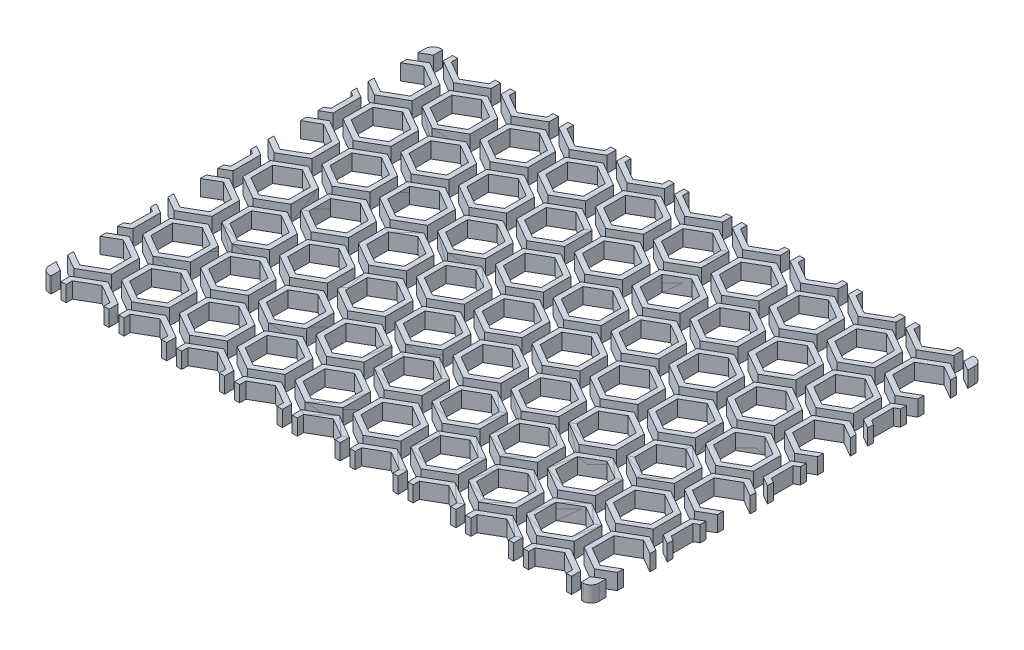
SolidWorks part; units mm, degrees
ref_plane "Front Plane" through (0, 0, 0) normal (0, 0, 1) x (1, 0, 0)
ref_plane "Top Plane" through (0, 0, 0) normal (0, 1, 0) x (1, 0, 0)
ref_plane "Right Plane" through (0, 0, 0) normal (1, 0, 0) x (0, 0, -1)
sketch "Sketch1" plane through (0, 0, 0) normal (0, 1, 0) x (1, 0, 0)
  line L0 (0, 7) -> (0, -23.7638) construction
  line L7 (0, 7) -> (-6.0622, 3.5)
  line L8 (-6.0622, 3.5) -> (-6.0622, -3.5)
  line L9 (-6.0622, -3.5) -> (0, -7)
  line L10 (0, -7) -> (6.0622, -3.5)
  line L11 (6.0622, -3.5) -> (6.0622, 3.5)
  line L12 (6.0622, 3.5) -> (0, 7)
  line L19 (13.3744, -9.1651) -> (7.3122, -5.6651)
  line L20 (7.3122, -5.6651) -> (1.25, -9.1651)
  line L21 (1.25, -9.1651) -> (1.25, -16.1651)
  line L22 (1.25, -16.1651) -> (7.3122, -19.6651)
  line L23 (7.3122, -19.6651) -> (13.3744, -16.1651)
  line L24 (13.3744, -16.1651) -> (13.3744, -9.1651)
  line L25 (14.62, 7) -> (8.5578, 3.5)
  line L26 (8.5578, -3.5) -> (14.62, -7)
  line L27 (8.5578, 3.5) -> (8.5578, -3.5)
  line L28 (20.6822, 3.5) -> (14.62, 7)
  line L29 (20.6822, -3.5) -> (20.6822, 3.5)
  line L30 (21.9322, -5.6651) -> (15.87, -9.1651)
  line L31 (27.9944, -9.1651) -> (21.9322, -5.6651)
  line L32 (27.9944, -16.1651) -> (27.9944, -9.1651)
  line L33 (21.9322, -19.6651) -> (27.9944, -16.1651)
  line L34 (15.87, -16.1651) -> (21.9322, -19.6651)
  line L35 (15.87, -9.1651) -> (15.87, -16.1651)
  line L36 (14.62, -7) -> (20.6822, -3.5)
  line L37 (29.24, 7) -> (23.1778, 3.5)
  line L38 (23.1778, -3.5) -> (29.24, -7)
  line L39 (23.1778, 3.5) -> (23.1778, -3.5)
  line L40 (35.3022, 3.5) -> (29.24, 7)
  line L41 (35.3022, -3.5) -> (35.3022, 3.5)
  line L42 (36.5522, -5.6651) -> (30.49, -9.1651)
  line L43 (42.6144, -9.1651) -> (36.5522, -5.6651)
  line L44 (42.6144, -16.1651) -> (42.6144, -9.1651)
  line L45 (36.5522, -19.6651) -> (42.6144, -16.1651)
  line L46 (30.49, -16.1651) -> (36.5522, -19.6651)
  line L47 (30.49, -9.1651) -> (30.49, -16.1651)
  line L48 (29.24, -7) -> (35.3022, -3.5)
  line L49 (43.86, 7) -> (37.7978, 3.5)
  line L50 (37.7978, -3.5) -> (43.86, -7)
  line L51 (37.7978, 3.5) -> (37.7978, -3.5)
  line L52 (49.9222, 3.5) -> (43.86, 7)
  line L53 (49.9222, -3.5) -> (49.9222, 3.5)
  line L54 (51.1722, -5.6651) -> (45.11, -9.1651)
  line L55 (57.2344, -9.1651) -> (51.1722, -5.6651)
  line L56 (57.2344, -16.1651) -> (57.2344, -9.1651)
  line L57 (51.1722, -19.6651) -> (57.2344, -16.1651)
  line L58 (45.11, -16.1651) -> (51.1722, -19.6651)
  line L59 (45.11, -9.1651) -> (45.11, -16.1651)
  line L60 (43.86, -7) -> (49.9222, -3.5)
  line L61 (14.62, -18.3301) -> (8.5578, -21.8301)
  line L62 (8.5578, -28.8301) -> (14.62, -32.3301)
  line L63 (8.5578, -21.8301) -> (8.5578, -28.8301)
  line L64 (20.6822, -21.8301) -> (14.62, -18.3301)
  line L65 (20.6822, -28.8301) -> (20.6822, -21.8301)
  line L66 (21.9322, -30.9952) -> (15.87, -34.4952)
  line L67 (27.9944, -34.4952) -> (21.9322, -30.9952)
  line L68 (27.9944, -41.4952) -> (27.9944, -34.4952)
  line L69 (21.9322, -44.9952) -> (27.9944, -41.4952)
  line L70 (15.87, -41.4952) -> (21.9322, -44.9952)
  line L71 (15.87, -34.4952) -> (15.87, -41.4952)
  line L72 (14.62, -32.3301) -> (20.6822, -28.8301)
  line L73 (29.24, -18.3301) -> (23.1778, -21.8301)
  line L74 (23.1778, -28.8301) -> (29.24, -32.3301)
  line L75 (23.1778, -21.8301) -> (23.1778, -28.8301)
  line L76 (35.3022, -21.8301) -> (29.24, -18.3301)
  line L77 (35.3022, -28.8301) -> (35.3022, -21.8301)
  line L78 (36.5522, -30.9952) -> (30.49, -34.4952)
  line L79 (42.6144, -34.4952) -> (36.5522, -30.9952)
  line L80 (42.6144, -41.4952) -> (42.6144, -34.4952)
  line L81 (36.5522, -44.9952) -> (42.6144, -41.4952)
  line L82 (30.49, -41.4952) -> (36.5522, -44.9952)
  line L83 (30.49, -34.4952) -> (30.49, -41.4952)
  line L84 (29.24, -32.3301) -> (35.3022, -28.8301)
  line L85 (43.86, -18.3301) -> (37.7978, -21.8301)
  line L86 (37.7978, -28.8301) -> (43.86, -32.3301)
  line L87 (37.7978, -21.8301) -> (37.7978, -28.8301)
  line L88 (49.9222, -21.8301) -> (43.86, -18.3301)
  line L89 (49.9222, -28.8301) -> (49.9222, -21.8301)
  line L90 (51.1722, -30.9952) -> (45.11, -34.4952)
  line L91 (57.2344, -34.4952) -> (51.1722, -30.9952)
  line L92 (57.2344, -41.4952) -> (57.2344, -34.4952)
  line L93 (51.1722, -44.9952) -> (57.2344, -41.4952)
  line L94 (45.11, -41.4952) -> (51.1722, -44.9952)
  line L95 (45.11, -34.4952) -> (45.11, -41.4952)
  line L96 (43.86, -32.3301) -> (49.9222, -28.8301)
  line L97 (14.62, -43.6603) -> (8.5578, -47.1603)
  line L98 (8.5578, -54.1603) -> (14.62, -57.6603)
  line L99 (8.5578, -47.1603) -> (8.5578, -54.1603)
  line L100 (20.6822, -47.1603) -> (14.62, -43.6603)
  line L101 (20.6822, -54.1603) -> (20.6822, -47.1603)
  line L102 (21.9322, -56.3253) -> (15.87, -59.8253)
  line L103 (27.9944, -59.8253) -> (21.9322, -56.3253)
  line L104 (27.9944, -66.8253) -> (27.9944, -59.8253)
  line L105 (21.9322, -70.3253) -> (27.9944, -66.8253)
  line L106 (15.87, -66.8253) -> (21.9322, -70.3253)
  line L107 (15.87, -59.8253) -> (15.87, -66.8253)
  line L108 (14.62, -57.6603) -> (20.6822, -54.1603)
  line L109 (29.24, -43.6603) -> (23.1778, -47.1603)
  line L110 (23.1778, -54.1603) -> (29.24, -57.6603)
  line L111 (23.1778, -47.1603) -> (23.1778, -54.1603)
  line L112 (35.3022, -47.1603) -> (29.24, -43.6603)
  line L113 (35.3022, -54.1603) -> (35.3022, -47.1603)
  line L114 (36.5522, -56.3253) -> (30.49, -59.8253)
  line L115 (42.6144, -59.8253) -> (36.5522, -56.3253)
  line L116 (42.6144, -66.8253) -> (42.6144, -59.8253)
  line L117 (36.5522, -70.3253) -> (42.6144, -66.8253)
  line L118 (30.49, -66.8253) -> (36.5522, -70.3253)
  line L119 (30.49, -59.8253) -> (30.49, -66.8253)
  line L120 (29.24, -57.6603) -> (35.3022, -54.1603)
  line L121 (43.86, -43.6603) -> (37.7978, -47.1603)
  line L122 (37.7978, -54.1603) -> (43.86, -57.6603)
  line L123 (37.7978, -47.1603) -> (37.7978, -54.1603)
  line L124 (49.9222, -47.1603) -> (43.86, -43.6603)
  line L125 (49.9222, -54.1603) -> (49.9222, -47.1603)
  line L126 (51.1722, -56.3253) -> (45.11, -59.8253)
  line L127 (57.2344, -59.8253) -> (51.1722, -56.3253)
  line L128 (57.2344, -66.8253) -> (57.2344, -59.8253)
  line L129 (51.1722, -70.3253) -> (57.2344, -66.8253)
  line L130 (45.11, -66.8253) -> (51.1722, -70.3253)
  line L131 (45.11, -59.8253) -> (45.11, -66.8253)
  line L132 (43.86, -57.6603) -> (49.9222, -54.1603)
  line L133 (0, -18.3301) -> (-6.0622, -21.8301)
  line L134 (-6.0622, -28.8301) -> (0, -32.3301)
  line L135 (-6.0622, -21.8301) -> (-6.0622, -28.8301)
  line L136 (6.0622, -21.8301) -> (0, -18.3301)
  line L137 (6.0622, -28.8301) -> (6.0622, -21.8301)
  line L138 (7.3122, -30.9952) -> (1.25, -34.4952)
  line L139 (13.3744, -34.4952) -> (7.3122, -30.9952)
  line L140 (13.3744, -41.4952) -> (13.3744, -34.4952)
  line L141 (7.3122, -44.9952) -> (13.3744, -41.4952)
  line L142 (1.25, -41.4952) -> (7.3122, -44.9952)
  line L143 (1.25, -34.4952) -> (1.25, -41.4952)
  line L144 (0, -32.3301) -> (6.0622, -28.8301)
  line L145 (0, -43.6603) -> (-6.0622, -47.1603)
  line L146 (-6.0622, -54.1603) -> (0, -57.6603)
  line L147 (-6.0622, -47.1603) -> (-6.0622, -54.1603)
  line L148 (6.0622, -47.1603) -> (0, -43.6603)
  line L149 (6.0622, -54.1603) -> (6.0622, -47.1603)
  line L150 (7.3122, -56.3253) -> (1.25, -59.8253)
  line L151 (13.3744, -59.8253) -> (7.3122, -56.3253)
  line L152 (13.3744, -66.8253) -> (13.3744, -59.8253)
  line L153 (7.3122, -70.3253) -> (13.3744, -66.8253)
  line L154 (1.25, -66.8253) -> (7.3122, -70.3253)
  line L155 (1.25, -59.8253) -> (1.25, -66.8253)
  line L156 (0, -57.6603) -> (6.0622, -54.1603)
  line L157 (-14.62, 7) -> (-20.6822, 3.5)
  line L158 (-8.5578, 3.5) -> (-14.62, 7)
  line L159 (-20.6822, 3.5) -> (-20.6822, -3.5)
  line L160 (-20.6822, -3.5) -> (-14.62, -7)
  line L161 (-14.62, -7) -> (-8.5578, -3.5)
  line L162 (-8.5578, -3.5) -> (-8.5578, 3.5)
  line L163 (-1.2456, -9.1651) -> (-7.3078, -5.6651)
  line L164 (-1.2456, -16.1651) -> (-1.2456, -9.1651)
  line L165 (-7.3078, -19.6651) -> (-1.2456, -16.1651)
  line L166 (-13.37, -16.1651) -> (-7.3078, -19.6651)
  line L167 (-13.37, -9.1651) -> (-13.37, -16.1651)
  line L168 (-7.3078, -5.6651) -> (-13.37, -9.1651)
  line L169 (-29.24, 7) -> (-35.3022, 3.5)
  line L170 (-23.1778, 3.5) -> (-29.24, 7)
  line L171 (-35.3022, 3.5) -> (-35.3022, -3.5)
  line L172 (-35.3022, -3.5) -> (-29.24, -7)
  line L173 (-29.24, -7) -> (-23.1778, -3.5)
  line L174 (-23.1778, -3.5) -> (-23.1778, 3.5)
  line L175 (-15.8656, -9.1651) -> (-21.9278, -5.6651)
  line L176 (-15.8656, -16.1651) -> (-15.8656, -9.1651)
  line L177 (-21.9278, -19.6651) -> (-15.8656, -16.1651)
  line L178 (-27.99, -16.1651) -> (-21.9278, -19.6651)
  line L179 (-27.99, -9.1651) -> (-27.99, -16.1651)
  line L180 (-21.9278, -5.6651) -> (-27.99, -9.1651)
  line L181 (-43.86, 7) -> (-49.9222, 3.5)
  line L182 (-37.7978, 3.5) -> (-43.86, 7)
  line L183 (-49.9222, 3.5) -> (-49.9222, -3.5)
  line L184 (-49.9222, -3.5) -> (-43.86, -7)
  line L185 (-43.86, -7) -> (-37.7978, -3.5)
  line L186 (-37.7978, -3.5) -> (-37.7978, 3.5)
  line L187 (-30.4856, -9.1651) -> (-36.5478, -5.6651)
  line L188 (-30.4856, -16.1651) -> (-30.4856, -9.1651)
  line L189 (-36.5478, -19.6651) -> (-30.4856, -16.1651)
  line L190 (-42.61, -16.1651) -> (-36.5478, -19.6651)
  line L191 (-42.61, -9.1651) -> (-42.61, -16.1651)
  line L192 (-36.5478, -5.6651) -> (-42.61, -9.1651)
  line L193 (-58.48, 7) -> (-64.5422, 3.5)
  line L194 (-52.4178, 3.5) -> (-58.48, 7)
  line L195 (-64.5422, 3.5) -> (-64.5422, -3.5)
  line L196 (-64.5422, -3.5) -> (-58.48, -7)
  line L197 (-58.48, -7) -> (-52.4178, -3.5)
  line L198 (-52.4178, -3.5) -> (-52.4178, 3.5)
  line L199 (-45.1056, -9.1651) -> (-51.1678, -5.6651)
  line L200 (-45.1056, -16.1651) -> (-45.1056, -9.1651)
  line L201 (-51.1678, -19.6651) -> (-45.1056, -16.1651)
  line L202 (-57.23, -16.1651) -> (-51.1678, -19.6651)
  line L203 (-57.23, -9.1651) -> (-57.23, -16.1651)
  line L204 (-51.1678, -5.6651) -> (-57.23, -9.1651)
  line L205 (-14.62, -18.33) -> (-20.6822, -21.83)
  line L206 (-8.5578, -21.83) -> (-14.62, -18.33)
  line L207 (-20.6822, -21.83) -> (-20.6822, -28.83)
  line L208 (-20.6822, -28.83) -> (-14.62, -32.33)
  line L209 (-14.62, -32.33) -> (-8.5578, -28.83)
  line L210 (-8.5578, -28.83) -> (-8.5578, -21.83)
  line L211 (-1.2456, -34.4951) -> (-7.3078, -30.9951)
  line L212 (-1.2456, -41.4951) -> (-1.2456, -34.4951)
  line L213 (-7.3078, -44.9951) -> (-1.2456, -41.4951)
  line L214 (-13.37, -41.4951) -> (-7.3078, -44.9951)
  line L215 (-13.37, -34.4951) -> (-13.37, -41.4951)
  line L216 (-7.3078, -30.9951) -> (-13.37, -34.4951)
  line L217 (-29.24, -18.33) -> (-35.3022, -21.83)
  line L218 (-23.1778, -21.83) -> (-29.24, -18.33)
  line L219 (-35.3022, -21.83) -> (-35.3022, -28.83)
  line L220 (-35.3022, -28.83) -> (-29.24, -32.33)
  line L221 (-29.24, -32.33) -> (-23.1778, -28.83)
  line L222 (-23.1778, -28.83) -> (-23.1778, -21.83)
  line L223 (-15.8656, -34.4951) -> (-21.9278, -30.9951)
  line L224 (-15.8656, -41.4951) -> (-15.8656, -34.4951)
  line L225 (-21.9278, -44.9951) -> (-15.8656, -41.4951)
  line L226 (-27.99, -41.4951) -> (-21.9278, -44.9951)
  line L227 (-27.99, -34.4951) -> (-27.99, -41.4951)
  line L228 (-21.9278, -30.9951) -> (-27.99, -34.4951)
  line L229 (-43.86, -18.33) -> (-49.9222, -21.83)
  line L230 (-37.7978, -21.83) -> (-43.86, -18.33)
  line L231 (-49.9222, -21.83) -> (-49.9222, -28.83)
  line L232 (-49.9222, -28.83) -> (-43.86, -32.33)
  line L233 (-43.86, -32.33) -> (-37.7978, -28.83)
  line L234 (-37.7978, -28.83) -> (-37.7978, -21.83)
  line L235 (-30.4856, -34.4951) -> (-36.5478, -30.9951)
  line L236 (-30.4856, -41.4951) -> (-30.4856, -34.4951)
  line L237 (-36.5478, -44.9951) -> (-30.4856, -41.4951)
  line L238 (-42.61, -41.4951) -> (-36.5478, -44.9951)
  line L239 (-42.61, -34.4951) -> (-42.61, -41.4951)
  line L240 (-36.5478, -30.9951) -> (-42.61, -34.4951)
  line L241 (-58.48, -18.33) -> (-64.5422, -21.83)
  line L242 (-52.4178, -21.83) -> (-58.48, -18.33)
  line L243 (-64.5422, -21.83) -> (-64.5422, -28.83)
  line L244 (-64.5422, -28.83) -> (-58.48, -32.33)
  line L245 (-58.48, -32.33) -> (-52.4178, -28.83)
  line L246 (-52.4178, -28.83) -> (-52.4178, -21.83)
  line L247 (-45.1056, -34.4951) -> (-51.1678, -30.9951)
  line L248 (-45.1056, -41.4951) -> (-45.1056, -34.4951)
  line L249 (-51.1678, -44.9951) -> (-45.1056, -41.4951)
  line L250 (-57.23, -41.4951) -> (-51.1678, -44.9951)
  line L251 (-57.23, -34.4951) -> (-57.23, -41.4951)
  line L252 (-51.1678, -30.9951) -> (-57.23, -34.4951)
  line L253 (-14.62, -43.66) -> (-20.6822, -47.16)
  line L254 (-8.5578, -47.16) -> (-14.62, -43.66)
  line L255 (-20.6822, -47.16) -> (-20.6822, -54.16)
  line L256 (-20.6822, -54.16) -> (-14.62, -57.66)
  line L257 (-14.62, -57.66) -> (-8.5578, -54.16)
  line L258 (-8.5578, -54.16) -> (-8.5578, -47.16)
  line L259 (-1.2456, -59.8251) -> (-7.3078, -56.3251)
  line L260 (-1.2456, -66.8251) -> (-1.2456, -59.8251)
  line L261 (-7.3078, -70.3251) -> (-1.2456, -66.8251)
  line L262 (-13.37, -66.8251) -> (-7.3078, -70.3251)
  line L263 (-13.37, -59.8251) -> (-13.37, -66.8251)
  line L264 (-7.3078, -56.3251) -> (-13.37, -59.8251)
  line L265 (-29.24, -43.66) -> (-35.3022, -47.16)
  line L266 (-23.1778, -47.16) -> (-29.24, -43.66)
  line L267 (-35.3022, -47.16) -> (-35.3022, -54.16)
  line L268 (-35.3022, -54.16) -> (-29.24, -57.66)
  line L269 (-29.24, -57.66) -> (-23.1778, -54.16)
  line L270 (-23.1778, -54.16) -> (-23.1778, -47.16)
  line L271 (-15.8656, -59.8251) -> (-21.9278, -56.3251)
  line L272 (-15.8656, -66.8251) -> (-15.8656, -59.8251)
  line L273 (-21.9278, -70.3251) -> (-15.8656, -66.8251)
  line L274 (-27.99, -66.8251) -> (-21.9278, -70.3251)
  line L275 (-27.99, -59.8251) -> (-27.99, -66.8251)
  line L276 (-21.9278, -56.3251) -> (-27.99, -59.8251)
  line L277 (-43.86, -43.66) -> (-49.9222, -47.16)
  line L278 (-37.7978, -47.16) -> (-43.86, -43.66)
  line L279 (-49.9222, -47.16) -> (-49.9222, -54.16)
  line L280 (-49.9222, -54.16) -> (-43.86, -57.66)
  line L281 (-43.86, -57.66) -> (-37.7978, -54.16)
  line L282 (-37.7978, -54.16) -> (-37.7978, -47.16)
  line L283 (-30.4856, -59.8251) -> (-36.5478, -56.3251)
  line L284 (-30.4856, -66.8251) -> (-30.4856, -59.8251)
  line L285 (-36.5478, -70.3251) -> (-30.4856, -66.8251)
  line L286 (-42.61, -66.8251) -> (-36.5478, -70.3251)
  line L287 (-42.61, -59.8251) -> (-42.61, -66.8251)
  line L288 (-36.5478, -56.3251) -> (-42.61, -59.8251)
  line L289 (-58.48, -43.66) -> (-64.5422, -47.16)
  line L290 (-52.4178, -47.16) -> (-58.48, -43.66)
  line L291 (-64.5422, -47.16) -> (-64.5422, -54.16)
  line L292 (-64.5422, -54.16) -> (-58.48, -57.66)
  line L293 (-58.48, -57.66) -> (-52.4178, -54.16)
  line L294 (-52.4178, -54.16) -> (-52.4178, -47.16)
  line L295 (-45.1056, -59.8251) -> (-51.1678, -56.3251)
  line L296 (-45.1056, -66.8251) -> (-45.1056, -59.8251)
  line L297 (-51.1678, -70.3251) -> (-45.1056, -66.8251)
  line L298 (-57.23, -66.8251) -> (-51.1678, -70.3251)
  line L299 (-57.23, -59.8251) -> (-57.23, -66.8251)
  line L300 (-51.1678, -56.3251) -> (-57.23, -59.8251)
  line L301 (0, -18.33) -> (-6.0622, -21.83)
  line L302 (6.0622, -21.83) -> (0, -18.33)
  line L303 (-6.0622, -21.83) -> (-6.0622, -28.83)
  line L304 (-6.0622, -28.83) -> (0, -32.33)
  line L305 (0, -32.33) -> (6.0622, -28.83)
  line L306 (6.0622, -28.83) -> (6.0622, -21.83)
  line L307 (13.3744, -34.4951) -> (7.3122, -30.9951)
  line L308 (13.3744, -41.4951) -> (13.3744, -34.4951)
  line L309 (7.3122, -44.9951) -> (13.3744, -41.4951)
  line L310 (1.25, -41.4951) -> (7.3122, -44.9951)
  line L311 (1.25, -34.4951) -> (1.25, -41.4951)
  line L312 (7.3122, -30.9951) -> (1.25, -34.4951)
  line L313 (0, -43.66) -> (-6.0622, -47.16)
  line L314 (6.0622, -47.16) -> (0, -43.66)
  line L315 (-6.0622, -47.16) -> (-6.0622, -54.16)
  line L316 (-6.0622, -54.16) -> (0, -57.66)
  line L317 (0, -57.66) -> (6.0622, -54.16)
  line L318 (6.0622, -54.16) -> (6.0622, -47.16)
  line L319 (13.3744, -59.8251) -> (7.3122, -56.3251)
  line L320 (13.3744, -66.8251) -> (13.3744, -59.8251)
  line L321 (7.3122, -70.3251) -> (13.3744, -66.8251)
  line L322 (1.25, -66.8251) -> (7.3122, -70.3251)
  line L323 (1.25, -59.8251) -> (1.25, -66.8251)
  line L324 (7.3122, -56.3251) -> (1.25, -59.8251)
  line L325 (14.62, 7) -> (8.5578, 3.5)
  line L326 (20.6822, 3.5) -> (14.62, 7)
  line L327 (8.5578, 3.5) -> (8.5578, -3.5)
  line L328 (8.5578, -3.5) -> (14.62, -7)
  line L329 (14.62, -7) -> (20.6822, -3.5)
  line L330 (20.6822, -3.5) -> (20.6822, 3.5)
  line L331 (27.9944, -9.1651) -> (21.9322, -5.6651)
  line L332 (27.9944, -16.1651) -> (27.9944, -9.1651)
  line L333 (21.9322, -19.6651) -> (27.9944, -16.1651)
  line L334 (15.87, -16.1651) -> (21.9322, -19.6651)
  line L335 (15.87, -9.1651) -> (15.87, -16.1651)
  line L336 (21.9322, -5.6651) -> (15.87, -9.1651)
  line L337 (29.24, 7) -> (23.1778, 3.5)
  line L338 (35.3022, 3.5) -> (29.24, 7)
  line L339 (23.1778, 3.5) -> (23.1778, -3.5)
  line L340 (23.1778, -3.5) -> (29.24, -7)
  line L341 (29.24, -7) -> (35.3022, -3.5)
  line L342 (35.3022, -3.5) -> (35.3022, 3.5)
  line L343 (42.6144, -9.1651) -> (36.5522, -5.6651)
  line L344 (42.6144, -16.1651) -> (42.6144, -9.1651)
  line L345 (36.5522, -19.6651) -> (42.6144, -16.1651)
  line L346 (30.49, -16.1651) -> (36.5522, -19.6651)
  line L347 (30.49, -9.1651) -> (30.49, -16.1651)
  line L348 (36.5522, -5.6651) -> (30.49, -9.1651)
  line L349 (43.86, 7) -> (37.7978, 3.5)
  line L350 (49.9222, 3.5) -> (43.86, 7)
  line L351 (37.7978, 3.5) -> (37.7978, -3.5)
  line L352 (37.7978, -3.5) -> (43.86, -7)
  line L353 (43.86, -7) -> (49.9222, -3.5)
  line L354 (49.9222, -3.5) -> (49.9222, 3.5)
  line L355 (57.2344, -9.1651) -> (51.1722, -5.6651)
  line L356 (57.2344, -16.1651) -> (57.2344, -9.1651)
  line L357 (51.1722, -19.6651) -> (57.2344, -16.1651)
  line L358 (45.11, -16.1651) -> (51.1722, -19.6651)
  line L359 (45.11, -9.1651) -> (45.11, -16.1651)
  line L360 (51.1722, -5.6651) -> (45.11, -9.1651)
  line L361 (14.62, 32.33) -> (8.5578, 28.83)
  line L362 (20.6822, 28.83) -> (14.62, 32.33)
  line L363 (8.5578, 28.83) -> (8.5578, 21.83)
  line L364 (8.5578, 21.83) -> (14.62, 18.33)
  line L365 (14.62, 18.33) -> (20.6822, 21.83)
  line L366 (20.6822, 21.83) -> (20.6822, 28.83)
  line L367 (27.9944, 16.1649) -> (21.9322, 19.6649)
  line L368 (27.9944, 9.1649) -> (27.9944, 16.1649)
  line L369 (21.9322, 5.6649) -> (27.9944, 9.1649)
  line L370 (15.87, 9.1649) -> (21.9322, 5.6649)
  line L371 (15.87, 16.1649) -> (15.87, 9.1649)
  line L372 (21.9322, 19.6649) -> (15.87, 16.1649)
  line L373 (29.24, 32.33) -> (23.1778, 28.83)
  line L374 (35.3022, 28.83) -> (29.24, 32.33)
  line L375 (23.1778, 28.83) -> (23.1778, 21.83)
  line L376 (23.1778, 21.83) -> (29.24, 18.33)
  line L377 (29.24, 18.33) -> (35.3022, 21.83)
  line L378 (35.3022, 21.83) -> (35.3022, 28.83)
  line L379 (42.6144, 16.1649) -> (36.5522, 19.6649)
  line L380 (42.6144, 9.1649) -> (42.6144, 16.1649)
  line L381 (36.5522, 5.6649) -> (42.6144, 9.1649)
  line L382 (30.49, 9.1649) -> (36.5522, 5.6649)
  line L383 (30.49, 16.1649) -> (30.49, 9.1649)
  line L384 (36.5522, 19.6649) -> (30.49, 16.1649)
  line L385 (43.86, 32.33) -> (37.7978, 28.83)
  line L386 (49.9222, 28.83) -> (43.86, 32.33)
  line L387 (37.7978, 28.83) -> (37.7978, 21.83)
  line L388 (37.7978, 21.83) -> (43.86, 18.33)
  line L389 (43.86, 18.33) -> (49.9222, 21.83)
  line L390 (49.9222, 21.83) -> (49.9222, 28.83)
  line L391 (57.2344, 16.1649) -> (51.1722, 19.6649)
  line L392 (57.2344, 9.1649) -> (57.2344, 16.1649)
  line L393 (51.1722, 5.6649) -> (57.2344, 9.1649)
  line L394 (45.11, 9.1649) -> (51.1722, 5.6649)
  line L395 (45.11, 16.1649) -> (45.11, 9.1649)
  line L396 (51.1722, 19.6649) -> (45.11, 16.1649)
  line L397 (14.62, 57.66) -> (8.5578, 54.16)
  line L398 (20.6822, 54.16) -> (14.62, 57.66)
  line L399 (8.5578, 54.16) -> (8.5578, 47.16)
  line L400 (8.5578, 47.16) -> (14.62, 43.66)
  line L401 (14.62, 43.66) -> (20.6822, 47.16)
  line L402 (20.6822, 47.16) -> (20.6822, 54.16)
  line L403 (27.9944, 41.4949) -> (21.9322, 44.9949)
  line L404 (27.9944, 34.4949) -> (27.9944, 41.4949)
  line L405 (21.9322, 30.9949) -> (27.9944, 34.4949)
  line L406 (15.87, 34.4949) -> (21.9322, 30.9949)
  line L407 (15.87, 41.4949) -> (15.87, 34.4949)
  line L408 (21.9322, 44.9949) -> (15.87, 41.4949)
  line L409 (29.24, 57.66) -> (23.1778, 54.16)
  line L410 (35.3022, 54.16) -> (29.24, 57.66)
  line L411 (23.1778, 54.16) -> (23.1778, 47.16)
  line L412 (23.1778, 47.16) -> (29.24, 43.66)
  line L413 (29.24, 43.66) -> (35.3022, 47.16)
  line L414 (35.3022, 47.16) -> (35.3022, 54.16)
  line L415 (42.6144, 41.4949) -> (36.5522, 44.9949)
  line L416 (42.6144, 34.4949) -> (42.6144, 41.4949)
  line L417 (36.5522, 30.9949) -> (42.6144, 34.4949)
  line L418 (30.49, 34.4949) -> (36.5522, 30.9949)
  line L419 (30.49, 41.4949) -> (30.49, 34.4949)
  line L420 (36.5522, 44.9949) -> (30.49, 41.4949)
  line L421 (43.86, 57.66) -> (37.7978, 54.16)
  line L422 (49.9222, 54.16) -> (43.86, 57.66)
  line L423 (37.7978, 54.16) -> (37.7978, 47.16)
  line L424 (37.7978, 47.16) -> (43.86, 43.66)
  line L425 (43.86, 43.66) -> (49.9222, 47.16)
  line L426 (49.9222, 47.16) -> (49.9222, 54.16)
  line L427 (57.2344, 41.4949) -> (51.1722, 44.9949)
  line L428 (57.2344, 34.4949) -> (57.2344, 41.4949)
  line L429 (51.1722, 30.9949) -> (57.2344, 34.4949)
  line L430 (45.11, 34.4949) -> (51.1722, 30.9949)
  line L431 (45.11, 41.4949) -> (45.11, 34.4949)
  line L432 (51.1722, 44.9949) -> (45.11, 41.4949)
  line L433 (14.62, 82.99) -> (8.5578, 79.49)
  line L434 (20.6822, 79.49) -> (14.62, 82.99)
  line L435 (8.5578, 79.49) -> (8.5578, 72.49)
  line L436 (8.5578, 72.49) -> (14.62, 68.99)
  line L437 (14.62, 68.99) -> (20.6822, 72.49)
  line L438 (20.6822, 72.49) -> (20.6822, 79.49)
  line L439 (27.9944, 66.8249) -> (21.9322, 70.3249)
  line L440 (27.9944, 59.8249) -> (27.9944, 66.8249)
  line L441 (21.9322, 56.3249) -> (27.9944, 59.8249)
  line L442 (15.87, 59.8249) -> (21.9322, 56.3249)
  line L443 (15.87, 66.8249) -> (15.87, 59.8249)
  line L444 (21.9322, 70.3249) -> (15.87, 66.8249)
  line L445 (29.24, 82.99) -> (23.1778, 79.49)
  line L446 (35.3022, 79.49) -> (29.24, 82.99)
  line L447 (23.1778, 79.49) -> (23.1778, 72.49)
  line L448 (23.1778, 72.49) -> (29.24, 68.99)
  line L449 (29.24, 68.99) -> (35.3022, 72.49)
  line L450 (35.3022, 72.49) -> (35.3022, 79.49)
  line L451 (42.6144, 66.8249) -> (36.5522, 70.3249)
  line L452 (42.6144, 59.8249) -> (42.6144, 66.8249)
  line L453 (36.5522, 56.3249) -> (42.6144, 59.8249)
  line L454 (30.49, 59.8249) -> (36.5522, 56.3249)
  line L455 (30.49, 66.8249) -> (30.49, 59.8249)
  line L456 (36.5522, 70.3249) -> (30.49, 66.8249)
  line L457 (43.86, 82.99) -> (37.7978, 79.49)
  line L458 (49.9222, 79.49) -> (43.86, 82.99)
  line L459 (37.7978, 79.49) -> (37.7978, 72.49)
  line L460 (37.7978, 72.49) -> (43.86, 68.99)
  line L461 (43.86, 68.99) -> (49.9222, 72.49)
  line L462 (49.9222, 72.49) -> (49.9222, 79.49)
  line L463 (57.2344, 66.8249) -> (51.1722, 70.3249)
  line L464 (57.2344, 59.8249) -> (57.2344, 66.8249)
  line L465 (51.1722, 56.3249) -> (57.2344, 59.8249)
  line L466 (45.11, 59.8249) -> (51.1722, 56.3249)
  line L467 (45.11, 66.8249) -> (45.11, 59.8249)
  line L468 (51.1722, 70.3249) -> (45.11, 66.8249)
  line L469 (0, 32.33) -> (-6.0622, 28.83)
  line L470 (6.0622, 28.83) -> (0, 32.33)
  line L471 (-6.0622, 28.83) -> (-6.0622, 21.83)
  line L472 (-6.0622, 21.83) -> (0, 18.33)
  line L473 (0, 18.33) -> (6.0622, 21.83)
  line L474 (6.0622, 21.83) -> (6.0622, 28.83)
  line L475 (13.3744, 16.1649) -> (7.3122, 19.6649)
  line L476 (13.3744, 9.1649) -> (13.3744, 16.1649)
  line L477 (7.3122, 5.6649) -> (13.3744, 9.1649)
  line L478 (1.25, 9.1649) -> (7.3122, 5.6649)
  line L479 (1.25, 16.1649) -> (1.25, 9.1649)
  line L480 (7.3122, 19.6649) -> (1.25, 16.1649)
  line L481 (0, 57.66) -> (-6.0622, 54.16)
  line L482 (6.0622, 54.16) -> (0, 57.66)
  line L483 (-6.0622, 54.16) -> (-6.0622, 47.16)
  line L484 (-6.0622, 47.16) -> (0, 43.66)
  line L485 (0, 43.66) -> (6.0622, 47.16)
  line L486 (6.0622, 47.16) -> (6.0622, 54.16)
  line L487 (13.3744, 41.4949) -> (7.3122, 44.9949)
  line L488 (13.3744, 34.4949) -> (13.3744, 41.4949)
  line L489 (7.3122, 30.9949) -> (13.3744, 34.4949)
  line L490 (1.25, 34.4949) -> (7.3122, 30.9949)
  line L491 (1.25, 41.4949) -> (1.25, 34.4949)
  line L492 (7.3122, 44.9949) -> (1.25, 41.4949)
  line L493 (0, 82.99) -> (-6.0622, 79.49)
  line L494 (6.0622, 79.49) -> (0, 82.99)
  line L495 (-6.0622, 79.49) -> (-6.0622, 72.49)
  line L496 (-6.0622, 72.49) -> (0, 68.99)
  line L497 (0, 68.99) -> (6.0622, 72.49)
  line L498 (6.0622, 72.49) -> (6.0622, 79.49)
  line L499 (13.3744, 66.8249) -> (7.3122, 70.3249)
  line L500 (13.3744, 59.8249) -> (13.3744, 66.8249)
  line L501 (7.3122, 56.3249) -> (13.3744, 59.8249)
  line L502 (1.25, 59.8249) -> (7.3122, 56.3249)
  line L503 (1.25, 66.8249) -> (1.25, 59.8249)
  line L504 (7.3122, 70.3249) -> (1.25, 66.8249)
  line L505 (-14.62, 7) -> (-20.6822, 3.5)
  line L506 (-8.5578, 3.5) -> (-14.62, 7)
  line L507 (-20.6822, 3.5) -> (-20.6822, -3.5)
  line L508 (-20.6822, -3.5) -> (-14.62, -7)
  line L509 (-14.62, -7) -> (-8.5578, -3.5)
  line L510 (-8.5578, -3.5) -> (-8.5578, 3.5)
  line L511 (-1.2456, -9.1651) -> (-7.3078, -5.6651)
  line L512 (-1.2456, -16.1651) -> (-1.2456, -9.1651)
  line L513 (-7.3078, -19.6651) -> (-1.2456, -16.1651)
  line L514 (-13.37, -16.1651) -> (-7.3078, -19.6651)
  line L515 (-13.37, -9.1651) -> (-13.37, -16.1651)
  line L516 (-7.3078, -5.6651) -> (-13.37, -9.1651)
  line L517 (-29.24, 7) -> (-35.3022, 3.5)
  line L518 (-23.1778, 3.5) -> (-29.24, 7)
  line L519 (-35.3022, 3.5) -> (-35.3022, -3.5)
  line L520 (-35.3022, -3.5) -> (-29.24, -7)
  line L521 (-29.24, -7) -> (-23.1778, -3.5)
  line L522 (-23.1778, -3.5) -> (-23.1778, 3.5)
  line L523 (-15.8656, -9.1651) -> (-21.9278, -5.6651)
  line L524 (-15.8656, -16.1651) -> (-15.8656, -9.1651)
  line L525 (-21.9278, -19.6651) -> (-15.8656, -16.1651)
  line L526 (-27.99, -16.1651) -> (-21.9278, -19.6651)
  line L527 (-27.99, -9.1651) -> (-27.99, -16.1651)
  line L528 (-21.9278, -5.6651) -> (-27.99, -9.1651)
  line L529 (-43.86, 7) -> (-49.9222, 3.5)
  line L530 (-37.7978, 3.5) -> (-43.86, 7)
  line L531 (-49.9222, 3.5) -> (-49.9222, -3.5)
  line L532 (-49.9222, -3.5) -> (-43.86, -7)
  line L533 (-43.86, -7) -> (-37.7978, -3.5)
  line L534 (-37.7978, -3.5) -> (-37.7978, 3.5)
  line L535 (-30.4856, -9.1651) -> (-36.5478, -5.6651)
  line L536 (-30.4856, -16.1651) -> (-30.4856, -9.1651)
  line L537 (-36.5478, -19.6651) -> (-30.4856, -16.1651)
  line L538 (-42.61, -16.1651) -> (-36.5478, -19.6651)
  line L539 (-42.61, -9.1651) -> (-42.61, -16.1651)
  line L540 (-36.5478, -5.6651) -> (-42.61, -9.1651)
  line L541 (-58.48, 7) -> (-64.5422, 3.5)
  line L542 (-52.4178, 3.5) -> (-58.48, 7)
  line L543 (-64.5422, 3.5) -> (-64.5422, -3.5)
  line L544 (-64.5422, -3.5) -> (-58.48, -7)
  line L545 (-58.48, -7) -> (-52.4178, -3.5)
  line L546 (-52.4178, -3.5) -> (-52.4178, 3.5)
  line L547 (-45.1056, -9.1651) -> (-51.1678, -5.6651)
  line L548 (-45.1056, -16.1651) -> (-45.1056, -9.1651)
  line L549 (-51.1678, -19.6651) -> (-45.1056, -16.1651)
  line L550 (-57.23, -16.1651) -> (-51.1678, -19.6651)
  line L551 (-57.23, -9.1651) -> (-57.23, -16.1651)
  line L552 (-51.1678, -5.6651) -> (-57.23, -9.1651)
  line L553 (-14.62, 32.33) -> (-20.6822, 28.83)
  line L554 (-8.5578, 28.83) -> (-14.62, 32.33)
  line L555 (-20.6822, 28.83) -> (-20.6822, 21.83)
  line L556 (-20.6822, 21.83) -> (-14.62, 18.33)
  line L557 (-14.62, 18.33) -> (-8.5578, 21.83)
  line L558 (-8.5578, 21.83) -> (-8.5578, 28.83)
  line L559 (-1.2456, 16.1649) -> (-7.3078, 19.6649)
  line L560 (-1.2456, 9.1649) -> (-1.2456, 16.1649)
  line L561 (-7.3078, 5.6649) -> (-1.2456, 9.1649)
  line L562 (-13.37, 9.1649) -> (-7.3078, 5.6649)
  line L563 (-13.37, 16.1649) -> (-13.37, 9.1649)
  line L564 (-7.3078, 19.6649) -> (-13.37, 16.1649)
  line L565 (-29.24, 32.33) -> (-35.3022, 28.83)
  line L566 (-23.1778, 28.83) -> (-29.24, 32.33)
  line L567 (-35.3022, 28.83) -> (-35.3022, 21.83)
  line L568 (-35.3022, 21.83) -> (-29.24, 18.33)
  line L569 (-29.24, 18.33) -> (-23.1778, 21.83)
  line L570 (-23.1778, 21.83) -> (-23.1778, 28.83)
  line L571 (-15.8656, 16.1649) -> (-21.9278, 19.6649)
  line L572 (-15.8656, 9.1649) -> (-15.8656, 16.1649)
  line L573 (-21.9278, 5.6649) -> (-15.8656, 9.1649)
  line L574 (-27.99, 9.1649) -> (-21.9278, 5.6649)
  line L575 (-27.99, 16.1649) -> (-27.99, 9.1649)
  line L576 (-21.9278, 19.6649) -> (-27.99, 16.1649)
  line L577 (-43.86, 32.33) -> (-49.9222, 28.83)
  line L578 (-37.7978, 28.83) -> (-43.86, 32.33)
  line L579 (-49.9222, 28.83) -> (-49.9222, 21.83)
  line L580 (-49.9222, 21.83) -> (-43.86, 18.33)
  line L581 (-43.86, 18.33) -> (-37.7978, 21.83)
  line L582 (-37.7978, 21.83) -> (-37.7978, 28.83)
  line L583 (-30.4856, 16.1649) -> (-36.5478, 19.6649)
  line L584 (-30.4856, 9.1649) -> (-30.4856, 16.1649)
  line L585 (-36.5478, 5.6649) -> (-30.4856, 9.1649)
  line L586 (-42.61, 9.1649) -> (-36.5478, 5.6649)
  line L587 (-42.61, 16.1649) -> (-42.61, 9.1649)
  line L588 (-36.5478, 19.6649) -> (-42.61, 16.1649)
  line L589 (-58.48, 32.33) -> (-64.5422, 28.83)
  line L590 (-52.4178, 28.83) -> (-58.48, 32.33)
  line L591 (-64.5422, 28.83) -> (-64.5422, 21.83)
  line L592 (-64.5422, 21.83) -> (-58.48, 18.33)
  line L593 (-58.48, 18.33) -> (-52.4178, 21.83)
  line L594 (-52.4178, 21.83) -> (-52.4178, 28.83)
  line L595 (-45.1056, 16.1649) -> (-51.1678, 19.6649)
  line L596 (-45.1056, 9.1649) -> (-45.1056, 16.1649)
  line L597 (-51.1678, 5.6649) -> (-45.1056, 9.1649)
  line L598 (-57.23, 9.1649) -> (-51.1678, 5.6649)
  line L599 (-57.23, 16.1649) -> (-57.23, 9.1649)
  line L600 (-51.1678, 19.6649) -> (-57.23, 16.1649)
  line L601 (-14.62, 57.66) -> (-20.6822, 54.16)
  line L602 (-8.5578, 54.16) -> (-14.62, 57.66)
  line L603 (-20.6822, 54.16) -> (-20.6822, 47.16)
  line L604 (-20.6822, 47.16) -> (-14.62, 43.66)
  line L605 (-14.62, 43.66) -> (-8.5578, 47.16)
  line L606 (-8.5578, 47.16) -> (-8.5578, 54.16)
  line L607 (-1.2456, 41.4949) -> (-7.3078, 44.9949)
  line L608 (-1.2456, 34.4949) -> (-1.2456, 41.4949)
  line L609 (-7.3078, 30.9949) -> (-1.2456, 34.4949)
  line L610 (-13.37, 34.4949) -> (-7.3078, 30.9949)
  line L611 (-13.37, 41.4949) -> (-13.37, 34.4949)
  line L612 (-7.3078, 44.9949) -> (-13.37, 41.4949)
  line L613 (-29.24, 57.66) -> (-35.3022, 54.16)
  line L614 (-23.1778, 54.16) -> (-29.24, 57.66)
  line L615 (-35.3022, 54.16) -> (-35.3022, 47.16)
  line L616 (-35.3022, 47.16) -> (-29.24, 43.66)
  line L617 (-29.24, 43.66) -> (-23.1778, 47.16)
  line L618 (-23.1778, 47.16) -> (-23.1778, 54.16)
  line L619 (-15.8656, 41.4949) -> (-21.9278, 44.9949)
  line L620 (-15.8656, 34.4949) -> (-15.8656, 41.4949)
  line L621 (-21.9278, 30.9949) -> (-15.8656, 34.4949)
  line L622 (-27.99, 34.4949) -> (-21.9278, 30.9949)
  line L623 (-27.99, 41.4949) -> (-27.99, 34.4949)
  line L624 (-21.9278, 44.9949) -> (-27.99, 41.4949)
  line L625 (-43.86, 57.66) -> (-49.9222, 54.16)
  line L626 (-37.7978, 54.16) -> (-43.86, 57.66)
  line L627 (-49.9222, 54.16) -> (-49.9222, 47.16)
  line L628 (-49.9222, 47.16) -> (-43.86, 43.66)
  line L629 (-43.86, 43.66) -> (-37.7978, 47.16)
  line L630 (-37.7978, 47.16) -> (-37.7978, 54.16)
  line L631 (-30.4856, 41.4949) -> (-36.5478, 44.9949)
  line L632 (-30.4856, 34.4949) -> (-30.4856, 41.4949)
  line L633 (-36.5478, 30.9949) -> (-30.4856, 34.4949)
  line L634 (-42.61, 34.4949) -> (-36.5478, 30.9949)
  line L635 (-42.61, 41.4949) -> (-42.61, 34.4949)
  line L636 (-36.5478, 44.9949) -> (-42.61, 41.4949)
  line L637 (-58.48, 57.66) -> (-64.5422, 54.16)
  line L638 (-52.4178, 54.16) -> (-58.48, 57.66)
  line L639 (-64.5422, 54.16) -> (-64.5422, 47.16)
  line L640 (-64.5422, 47.16) -> (-58.48, 43.66)
  line L641 (-58.48, 43.66) -> (-52.4178, 47.16)
  line L642 (-52.4178, 47.16) -> (-52.4178, 54.16)
  line L643 (-45.1056, 41.4949) -> (-51.1678, 44.9949)
  line L644 (-45.1056, 34.4949) -> (-45.1056, 41.4949)
  line L645 (-51.1678, 30.9949) -> (-45.1056, 34.4949)
  line L646 (-57.23, 34.4949) -> (-51.1678, 30.9949)
  line L647 (-57.23, 41.4949) -> (-57.23, 34.4949)
  line L648 (-51.1678, 44.9949) -> (-57.23, 41.4949)
  line L649 (-14.62, 82.99) -> (-20.6822, 79.49)
  line L650 (-8.5578, 79.49) -> (-14.62, 82.99)
  line L651 (-20.6822, 79.49) -> (-20.6822, 72.49)
  line L652 (-20.6822, 72.49) -> (-14.62, 68.99)
  line L653 (-14.62, 68.99) -> (-8.5578, 72.49)
  line L654 (-8.5578, 72.49) -> (-8.5578, 79.49)
  line L655 (-1.2456, 66.8249) -> (-7.3078, 70.3249)
  line L656 (-1.2456, 59.8249) -> (-1.2456, 66.8249)
  line L657 (-7.3078, 56.3249) -> (-1.2456, 59.8249)
  line L658 (-13.37, 59.8249) -> (-7.3078, 56.3249)
  line L659 (-13.37, 66.8249) -> (-13.37, 59.8249)
  line L660 (-7.3078, 70.3249) -> (-13.37, 66.8249)
  line L661 (-29.24, 82.99) -> (-35.3022, 79.49)
  line L662 (-23.1778, 79.49) -> (-29.24, 82.99)
  line L663 (-35.3022, 79.49) -> (-35.3022, 72.49)
  line L664 (-35.3022, 72.49) -> (-29.24, 68.99)
  line L665 (-29.24, 68.99) -> (-23.1778, 72.49)
  line L666 (-23.1778, 72.49) -> (-23.1778, 79.49)
  line L667 (-15.8656, 66.8249) -> (-21.9278, 70.3249)
  line L668 (-15.8656, 59.8249) -> (-15.8656, 66.8249)
  line L669 (-21.9278, 56.3249) -> (-15.8656, 59.8249)
  line L670 (-27.99, 59.8249) -> (-21.9278, 56.3249)
  line L671 (-27.99, 66.8249) -> (-27.99, 59.8249)
  line L672 (-21.9278, 70.3249) -> (-27.99, 66.8249)
  line L673 (-43.86, 82.99) -> (-49.9222, 79.49)
  line L674 (-37.7978, 79.49) -> (-43.86, 82.99)
  line L675 (-49.9222, 79.49) -> (-49.9222, 72.49)
  line L676 (-49.9222, 72.49) -> (-43.86, 68.99)
  line L677 (-43.86, 68.99) -> (-37.7978, 72.49)
  line L678 (-37.7978, 72.49) -> (-37.7978, 79.49)
  line L679 (-30.4856, 66.8249) -> (-36.5478, 70.3249)
  line L680 (-30.4856, 59.8249) -> (-30.4856, 66.8249)
  line L681 (-36.5478, 56.3249) -> (-30.4856, 59.8249)
  line L682 (-42.61, 59.8249) -> (-36.5478, 56.3249)
  line L683 (-42.61, 66.8249) -> (-42.61, 59.8249)
  line L684 (-36.5478, 70.3249) -> (-42.61, 66.8249)
  line L685 (-58.48, 82.99) -> (-64.5422, 79.49)
  line L686 (-52.4178, 79.49) -> (-58.48, 82.99)
  line L687 (-64.5422, 79.49) -> (-64.5422, 72.49)
  line L688 (-64.5422, 72.49) -> (-58.48, 68.99)
  line L689 (-58.48, 68.99) -> (-52.4178, 72.49)
  line L690 (-52.4178, 72.49) -> (-52.4178, 79.49)
  line L691 (-45.1056, 66.8249) -> (-51.1678, 70.3249)
  line L692 (-45.1056, 59.8249) -> (-45.1056, 66.8249)
  line L693 (-51.1678, 56.3249) -> (-45.1056, 59.8249)
  line L694 (-57.23, 59.8249) -> (-51.1678, 56.3249)
  line L695 (-57.23, 66.8249) -> (-57.23, 59.8249)
  line L696 (-51.1678, 70.3249) -> (-57.23, 66.8249)
  line L697 (0, 32.33) -> (-6.0622, 28.83)
  line L698 (6.0622, 28.83) -> (0, 32.33)
  line L699 (-6.0622, 28.83) -> (-6.0622, 21.83)
  line L700 (-6.0622, 21.83) -> (0, 18.33)
  line L701 (0, 18.33) -> (6.0622, 21.83)
  line L702 (6.0622, 21.83) -> (6.0622, 28.83)
  line L703 (13.3744, 16.1649) -> (7.3122, 19.6649)
  line L704 (13.3744, 9.1649) -> (13.3744, 16.1649)
  line L705 (7.3122, 5.6649) -> (13.3744, 9.1649)
  line L706 (1.25, 9.1649) -> (7.3122, 5.6649)
  line L707 (1.25, 16.1649) -> (1.25, 9.1649)
  line L708 (7.3122, 19.6649) -> (1.25, 16.1649)
  line L709 (0, 57.66) -> (-6.0622, 54.16)
  line L710 (6.0622, 54.16) -> (0, 57.66)
  line L711 (-6.0622, 54.16) -> (-6.0622, 47.16)
  line L712 (-6.0622, 47.16) -> (0, 43.66)
  line L713 (0, 43.66) -> (6.0622, 47.16)
  line L714 (6.0622, 47.16) -> (6.0622, 54.16)
  line L715 (13.3744, 41.4949) -> (7.3122, 44.9949)
  line L716 (13.3744, 34.4949) -> (13.3744, 41.4949)
  line L717 (7.3122, 30.9949) -> (13.3744, 34.4949)
  line L718 (1.25, 34.4949) -> (7.3122, 30.9949)
  line L719 (1.25, 41.4949) -> (1.25, 34.4949)
  line L720 (7.3122, 44.9949) -> (1.25, 41.4949)
  line L721 (0, 82.99) -> (-6.0622, 79.49)
  line L722 (6.0622, 79.49) -> (0, 82.99)
  line L723 (-6.0622, 79.49) -> (-6.0622, 72.49)
  line L724 (-6.0622, 72.49) -> (0, 68.99)
  line L725 (0, 68.99) -> (6.0622, 72.49)
  line L726 (6.0622, 72.49) -> (6.0622, 79.49)
  line L727 (13.3744, 66.8249) -> (7.3122, 70.3249)
  line L728 (13.3744, 59.8249) -> (13.3744, 66.8249)
  line L729 (7.3122, 56.3249) -> (13.3744, 59.8249)
  line L730 (1.25, 59.8249) -> (7.3122, 56.3249)
  line L731 (1.25, 66.8249) -> (1.25, 59.8249)
  line L732 (7.3122, 70.3249) -> (1.25, 66.8249)
  line L733 (14.62, -7) -> (20.6822, -3.5)
  line L734 (20.6822, -3.5) -> (20.6822, 3.5)
  line L735 (20.6822, 3.5) -> (14.62, 7)
  line L736 (14.62, 7) -> (8.5578, 3.5)
  line L737 (8.5578, 3.5) -> (8.5578, -3.5)
  line L738 (8.5578, -3.5) -> (14.62, -7)
  line L739 (21.9322, -5.6651) -> (15.87, -9.1651)
  line L740 (15.87, -9.1651) -> (15.87, -16.1651)
  line L741 (15.87, -16.1651) -> (21.9322, -19.6651)
  line L742 (21.9322, -19.6651) -> (27.9944, -16.1651)
  line L743 (27.9944, -16.1651) -> (27.9944, -9.1651)
  line L744 (27.9944, -9.1651) -> (21.9322, -5.6651)
  line L745 (29.24, -7) -> (35.3022, -3.5)
  line L746 (35.3022, -3.5) -> (35.3022, 3.5)
  line L747 (35.3022, 3.5) -> (29.24, 7)
  line L748 (29.24, 7) -> (23.1778, 3.5)
  line L749 (23.1778, 3.5) -> (23.1778, -3.5)
  line L750 (23.1778, -3.5) -> (29.24, -7)
  line L751 (36.5522, -5.6651) -> (30.49, -9.1651)
  line L752 (30.49, -9.1651) -> (30.49, -16.1651)
  line L753 (30.49, -16.1651) -> (36.5522, -19.6651)
  line L754 (36.5522, -19.6651) -> (42.6144, -16.1651)
  line L755 (42.6144, -16.1651) -> (42.6144, -9.1651)
  line L756 (42.6144, -9.1651) -> (36.5522, -5.6651)
  line L757 (43.86, -7) -> (49.9222, -3.5)
  line L758 (49.9222, -3.5) -> (49.9222, 3.5)
  line L759 (49.9222, 3.5) -> (43.86, 7)
  line L760 (43.86, 7) -> (37.7978, 3.5)
  line L761 (37.7978, 3.5) -> (37.7978, -3.5)
  line L762 (37.7978, -3.5) -> (43.86, -7)
  line L763 (51.1722, -5.6651) -> (45.11, -9.1651)
  line L764 (45.11, -9.1651) -> (45.11, -16.1651)
  line L765 (45.11, -16.1651) -> (51.1722, -19.6651)
  line L766 (51.1722, -19.6651) -> (57.2344, -16.1651)
  line L767 (57.2344, -16.1651) -> (57.2344, -9.1651)
  line L768 (57.2344, -9.1651) -> (51.1722, -5.6651)
  line L769 (58.48, -7) -> (64.5422, -3.5)
  line L770 (64.5422, -3.5) -> (64.5422, 3.5)
  line L771 (64.5422, 3.5) -> (58.48, 7)
  line L772 (58.48, 7) -> (52.4178, 3.5)
  line L773 (52.4178, 3.5) -> (52.4178, -3.5)
  line L774 (52.4178, -3.5) -> (58.48, -7)
  line L775 (65.7922, -5.6651) -> (59.73, -9.1651)
  line L776 (59.73, -9.1651) -> (59.73, -16.1651)
  line L777 (59.73, -16.1651) -> (65.7922, -19.6651)
  line L778 (65.7922, -19.6651) -> (71.8544, -16.1651)
  line L779 (71.8544, -16.1651) -> (71.8544, -9.1651)
  line L780 (71.8544, -9.1651) -> (65.7922, -5.6651)
  line L781 (73.1, -7) -> (79.1622, -3.5)
  line L782 (79.1622, -3.5) -> (79.1622, 3.5)
  line L783 (79.1622, 3.5) -> (73.1, 7)
  line L784 (73.1, 7) -> (67.0378, 3.5)
  line L785 (67.0378, 3.5) -> (67.0378, -3.5)
  line L786 (67.0378, -3.5) -> (73.1, -7)
  line L787 (80.4122, -5.6651) -> (74.35, -9.1651)
  line L788 (74.35, -9.1651) -> (74.35, -16.1651)
  line L789 (74.35, -16.1651) -> (80.4122, -19.6651)
  line L790 (80.4122, -19.6651) -> (86.4744, -16.1651)
  line L791 (86.4744, -16.1651) -> (86.4744, -9.1651)
  line L792 (86.4744, -9.1651) -> (80.4122, -5.6651)
  line L793 (87.72, -7) -> (93.7822, -3.5)
  line L794 (93.7822, -3.5) -> (93.7822, 3.5)
  line L795 (93.7822, 3.5) -> (87.72, 7)
  line L796 (87.72, 7) -> (81.6578, 3.5)
  line L797 (81.6578, 3.5) -> (81.6578, -3.5)
  line L798 (81.6578, -3.5) -> (87.72, -7)
  line L799 (95.0322, -5.6651) -> (88.97, -9.1651)
  line L800 (88.97, -9.1651) -> (88.97, -16.1651)
  line L801 (88.97, -16.1651) -> (95.0322, -19.6651)
  line L802 (95.0322, -19.6651) -> (101.0944, -16.1651)
  line L803 (101.0944, -16.1651) -> (101.0944, -9.1651)
  line L804 (101.0944, -9.1651) -> (95.0322, -5.6651)
  line L805 (14.62, 18.33) -> (20.6822, 21.83)
  line L806 (20.6822, 21.83) -> (20.6822, 28.83)
  line L807 (20.6822, 28.83) -> (14.62, 32.33)
  line L808 (14.62, 32.33) -> (8.5578, 28.83)
  line L809 (8.5578, 28.83) -> (8.5578, 21.83)
  line L810 (8.5578, 21.83) -> (14.62, 18.33)
  line L811 (21.9322, 19.6649) -> (15.87, 16.1649)
  line L812 (15.87, 16.1649) -> (15.87, 9.1649)
  line L813 (15.87, 9.1649) -> (21.9322, 5.6649)
  line L814 (21.9322, 5.6649) -> (27.9944, 9.1649)
  line L815 (27.9944, 9.1649) -> (27.9944, 16.1649)
  line L816 (27.9944, 16.1649) -> (21.9322, 19.6649)
  line L817 (29.24, 18.33) -> (35.3022, 21.83)
  line L818 (35.3022, 21.83) -> (35.3022, 28.83)
  line L819 (35.3022, 28.83) -> (29.24, 32.33)
  line L820 (29.24, 32.33) -> (23.1778, 28.83)
  line L821 (23.1778, 28.83) -> (23.1778, 21.83)
  line L822 (23.1778, 21.83) -> (29.24, 18.33)
  line L823 (36.5522, 19.6649) -> (30.49, 16.1649)
  line L824 (30.49, 16.1649) -> (30.49, 9.1649)
  line L825 (30.49, 9.1649) -> (36.5522, 5.6649)
  line L826 (36.5522, 5.6649) -> (42.6144, 9.1649)
  line L827 (42.6144, 9.1649) -> (42.6144, 16.1649)
  line L828 (42.6144, 16.1649) -> (36.5522, 19.6649)
  line L829 (43.86, 18.33) -> (49.9222, 21.83)
  line L830 (49.9222, 21.83) -> (49.9222, 28.83)
  line L831 (49.9222, 28.83) -> (43.86, 32.33)
  line L832 (43.86, 32.33) -> (37.7978, 28.83)
  line L833 (37.7978, 28.83) -> (37.7978, 21.83)
  line L834 (37.7978, 21.83) -> (43.86, 18.33)
  line L835 (51.1722, 19.6649) -> (45.11, 16.1649)
  line L836 (45.11, 16.1649) -> (45.11, 9.1649)
  line L837 (45.11, 9.1649) -> (51.1722, 5.6649)
  line L838 (51.1722, 5.6649) -> (57.2344, 9.1649)
  line L839 (57.2344, 9.1649) -> (57.2344, 16.1649)
  line L840 (57.2344, 16.1649) -> (51.1722, 19.6649)
  line L841 (58.48, 18.33) -> (64.5422, 21.83)
  line L842 (64.5422, 21.83) -> (64.5422, 28.83)
  line L843 (64.5422, 28.83) -> (58.48, 32.33)
  line L844 (58.48, 32.33) -> (52.4178, 28.83)
  line L845 (52.4178, 28.83) -> (52.4178, 21.83)
  line L846 (52.4178, 21.83) -> (58.48, 18.33)
  line L847 (65.7922, 19.6649) -> (59.73, 16.1649)
  line L848 (59.73, 16.1649) -> (59.73, 9.1649)
  line L849 (59.73, 9.1649) -> (65.7922, 5.6649)
  line L850 (65.7922, 5.6649) -> (71.8544, 9.1649)
  line L851 (71.8544, 9.1649) -> (71.8544, 16.1649)
  line L852 (71.8544, 16.1649) -> (65.7922, 19.6649)
  line L853 (73.1, 18.33) -> (79.1622, 21.83)
  line L854 (79.1622, 21.83) -> (79.1622, 28.83)
  line L855 (79.1622, 28.83) -> (73.1, 32.33)
  line L856 (73.1, 32.33) -> (67.0378, 28.83)
  line L857 (67.0378, 28.83) -> (67.0378, 21.83)
  line L858 (67.0378, 21.83) -> (73.1, 18.33)
  line L859 (80.4122, 19.6649) -> (74.35, 16.1649)
  line L860 (74.35, 16.1649) -> (74.35, 9.1649)
  line L861 (74.35, 9.1649) -> (80.4122, 5.6649)
  line L862 (80.4122, 5.6649) -> (86.4744, 9.1649)
  line L863 (86.4744, 9.1649) -> (86.4744, 16.1649)
  line L864 (86.4744, 16.1649) -> (80.4122, 19.6649)
  line L865 (87.72, 18.33) -> (93.7822, 21.83)
  line L866 (93.7822, 21.83) -> (93.7822, 28.83)
  line L867 (93.7822, 28.83) -> (87.72, 32.33)
  line L868 (87.72, 32.33) -> (81.6578, 28.83)
  line L869 (81.6578, 28.83) -> (81.6578, 21.83)
  line L870 (81.6578, 21.83) -> (87.72, 18.33)
  line L871 (95.0322, 19.6649) -> (88.97, 16.1649)
  line L872 (88.97, 16.1649) -> (88.97, 9.1649)
  line L873 (88.97, 9.1649) -> (95.0322, 5.6649)
  line L874 (95.0322, 5.6649) -> (101.0944, 9.1649)
  line L875 (101.0944, 9.1649) -> (101.0944, 16.1649)
  line L876 (101.0944, 16.1649) -> (95.0322, 19.6649)
  line L877 (14.62, 43.66) -> (20.6822, 47.16)
  line L878 (20.6822, 47.16) -> (20.6822, 54.16)
  line L879 (20.6822, 54.16) -> (14.62, 57.66)
  line L880 (14.62, 57.66) -> (8.5578, 54.16)
  line L881 (8.5578, 54.16) -> (8.5578, 47.16)
  line L882 (8.5578, 47.16) -> (14.62, 43.66)
  line L883 (21.9322, 44.9949) -> (15.87, 41.4949)
  line L884 (15.87, 41.4949) -> (15.87, 34.4949)
  line L885 (15.87, 34.4949) -> (21.9322, 30.9949)
  line L886 (21.9322, 30.9949) -> (27.9944, 34.4949)
  line L887 (27.9944, 34.4949) -> (27.9944, 41.4949)
  line L888 (27.9944, 41.4949) -> (21.9322, 44.9949)
  line L889 (29.24, 43.66) -> (35.3022, 47.16)
  line L890 (35.3022, 47.16) -> (35.3022, 54.16)
  line L891 (35.3022, 54.16) -> (29.24, 57.66)
  line L892 (29.24, 57.66) -> (23.1778, 54.16)
  line L893 (23.1778, 54.16) -> (23.1778, 47.16)
  line L894 (23.1778, 47.16) -> (29.24, 43.66)
  line L895 (36.5522, 44.9949) -> (30.49, 41.4949)
  line L896 (30.49, 41.4949) -> (30.49, 34.4949)
  line L897 (30.49, 34.4949) -> (36.5522, 30.9949)
  line L898 (36.5522, 30.9949) -> (42.6144, 34.4949)
  line L899 (42.6144, 34.4949) -> (42.6144, 41.4949)
  line L900 (42.6144, 41.4949) -> (36.5522, 44.9949)
  line L901 (43.86, 43.66) -> (49.9222, 47.16)
  line L902 (49.9222, 47.16) -> (49.9222, 54.16)
  line L903 (49.9222, 54.16) -> (43.86, 57.66)
  line L904 (43.86, 57.66) -> (37.7978, 54.16)
  line L905 (37.7978, 54.16) -> (37.7978, 47.16)
  line L906 (37.7978, 47.16) -> (43.86, 43.66)
  line L907 (51.1722, 44.9949) -> (45.11, 41.4949)
  line L908 (45.11, 41.4949) -> (45.11, 34.4949)
  line L909 (45.11, 34.4949) -> (51.1722, 30.9949)
  line L910 (51.1722, 30.9949) -> (57.2344, 34.4949)
  line L911 (57.2344, 34.4949) -> (57.2344, 41.4949)
  line L912 (57.2344, 41.4949) -> (51.1722, 44.9949)
  line L913 (58.48, 43.66) -> (64.5422, 47.16)
  line L914 (64.5422, 47.16) -> (64.5422, 54.16)
  line L915 (64.5422, 54.16) -> (58.48, 57.66)
  line L916 (58.48, 57.66) -> (52.4178, 54.16)
  line L917 (52.4178, 54.16) -> (52.4178, 47.16)
  line L918 (52.4178, 47.16) -> (58.48, 43.66)
  line L919 (65.7922, 44.9949) -> (59.73, 41.4949)
  line L920 (59.73, 41.4949) -> (59.73, 34.4949)
  line L921 (59.73, 34.4949) -> (65.7922, 30.9949)
  line L922 (65.7922, 30.9949) -> (71.8544, 34.4949)
  line L923 (71.8544, 34.4949) -> (71.8544, 41.4949)
  line L924 (71.8544, 41.4949) -> (65.7922, 44.9949)
  line L925 (73.1, 43.66) -> (79.1622, 47.16)
  line L926 (79.1622, 47.16) -> (79.1622, 54.16)
  line L927 (79.1622, 54.16) -> (73.1, 57.66)
  line L928 (73.1, 57.66) -> (67.0378, 54.16)
  line L929 (67.0378, 54.16) -> (67.0378, 47.16)
  line L930 (67.0378, 47.16) -> (73.1, 43.66)
  line L931 (80.4122, 44.9949) -> (74.35, 41.4949)
  line L932 (74.35, 41.4949) -> (74.35, 34.4949)
  line L933 (74.35, 34.4949) -> (80.4122, 30.9949)
  line L934 (80.4122, 30.9949) -> (86.4744, 34.4949)
  line L935 (86.4744, 34.4949) -> (86.4744, 41.4949)
  line L936 (86.4744, 41.4949) -> (80.4122, 44.9949)
  line L937 (87.72, 43.66) -> (93.7822, 47.16)
  line L938 (93.7822, 47.16) -> (93.7822, 54.16)
  line L939 (93.7822, 54.16) -> (87.72, 57.66)
  line L940 (87.72, 57.66) -> (81.6578, 54.16)
  line L941 (81.6578, 54.16) -> (81.6578, 47.16)
  line L942 (81.6578, 47.16) -> (87.72, 43.66)
  line L943 (95.0322, 44.9949) -> (88.97, 41.4949)
  line L944 (88.97, 41.4949) -> (88.97, 34.4949)
  line L945 (88.97, 34.4949) -> (95.0322, 30.9949)
  line L946 (95.0322, 30.9949) -> (101.0944, 34.4949)
  line L947 (101.0944, 34.4949) -> (101.0944, 41.4949)
  line L948 (101.0944, 41.4949) -> (95.0322, 44.9949)
  line L949 (14.62, 68.99) -> (20.6822, 72.49)
  line L950 (20.6822, 72.49) -> (20.6822, 79.49)
  line L951 (20.6822, 79.49) -> (14.62, 82.99)
  line L952 (14.62, 82.99) -> (8.5578, 79.49)
  line L953 (8.5578, 79.49) -> (8.5578, 72.49)
  line L954 (8.5578, 72.49) -> (14.62, 68.99)
  line L955 (21.9322, 70.3249) -> (15.87, 66.8249)
  line L956 (15.87, 66.8249) -> (15.87, 59.8249)
  line L957 (15.87, 59.8249) -> (21.9322, 56.3249)
  line L958 (21.9322, 56.3249) -> (27.9944, 59.8249)
  line L959 (27.9944, 59.8249) -> (27.9944, 66.8249)
  line L960 (27.9944, 66.8249) -> (21.9322, 70.3249)
  line L961 (29.24, 68.99) -> (35.3022, 72.49)
  line L962 (35.3022, 72.49) -> (35.3022, 79.49)
  line L963 (35.3022, 79.49) -> (29.24, 82.99)
  line L964 (29.24, 82.99) -> (23.1778, 79.49)
  line L965 (23.1778, 79.49) -> (23.1778, 72.49)
  line L966 (23.1778, 72.49) -> (29.24, 68.99)
  line L967 (36.5522, 70.3249) -> (30.49, 66.8249)
  line L968 (30.49, 66.8249) -> (30.49, 59.8249)
  line L969 (30.49, 59.8249) -> (36.5522, 56.3249)
  line L970 (36.5522, 56.3249) -> (42.6144, 59.8249)
  line L971 (42.6144, 59.8249) -> (42.6144, 66.8249)
  line L972 (42.6144, 66.8249) -> (36.5522, 70.3249)
  line L973 (43.86, 68.99) -> (49.9222, 72.49)
  line L974 (49.9222, 72.49) -> (49.9222, 79.49)
  line L975 (49.9222, 79.49) -> (43.86, 82.99)
  line L976 (43.86, 82.99) -> (37.7978, 79.49)
  line L977 (37.7978, 79.49) -> (37.7978, 72.49)
  line L978 (37.7978, 72.49) -> (43.86, 68.99)
  line L979 (51.1722, 70.3249) -> (45.11, 66.8249)
  line L980 (45.11, 66.8249) -> (45.11, 59.8249)
  line L981 (45.11, 59.8249) -> (51.1722, 56.3249)
  line L982 (51.1722, 56.3249) -> (57.2344, 59.8249)
  line L983 (57.2344, 59.8249) -> (57.2344, 66.8249)
  line L984 (57.2344, 66.8249) -> (51.1722, 70.3249)
  line L985 (58.48, 68.99) -> (64.5422, 72.49)
  line L986 (64.5422, 72.49) -> (64.5422, 79.49)
  line L987 (64.5422, 79.49) -> (58.48, 82.99)
  line L988 (58.48, 82.99) -> (52.4178, 79.49)
  line L989 (52.4178, 79.49) -> (52.4178, 72.49)
  line L990 (52.4178, 72.49) -> (58.48, 68.99)
  line L991 (65.7922, 70.3249) -> (59.73, 66.8249)
  line L992 (59.73, 66.8249) -> (59.73, 59.8249)
  line L993 (59.73, 59.8249) -> (65.7922, 56.3249)
  line L994 (65.7922, 56.3249) -> (71.8544, 59.8249)
  line L995 (71.8544, 59.8249) -> (71.8544, 66.8249)
  line L996 (71.8544, 66.8249) -> (65.7922, 70.3249)
  line L997 (73.1, 68.99) -> (79.1622, 72.49)
  line L998 (79.1622, 72.49) -> (79.1622, 79.49)
  line L999 (79.1622, 79.49) -> (73.1, 82.99)
  line L1000 (73.1, 82.99) -> (67.0378, 79.49)
  line L1001 (67.0378, 79.49) -> (67.0378, 72.49)
  line L1002 (67.0378, 72.49) -> (73.1, 68.99)
  line L1003 (80.4122, 70.3249) -> (74.35, 66.8249)
  line L1004 (74.35, 66.8249) -> (74.35, 59.8249)
  line L1005 (74.35, 59.8249) -> (80.4122, 56.3249)
  line L1006 (80.4122, 56.3249) -> (86.4744, 59.8249)
  line L1007 (86.4744, 59.8249) -> (86.4744, 66.8249)
  line L1008 (86.4744, 66.8249) -> (80.4122, 70.3249)
  line L1009 (87.72, 68.99) -> (93.7822, 72.49)
  line L1010 (93.7822, 72.49) -> (93.7822, 79.49)
  line L1011 (93.7822, 79.49) -> (87.72, 82.99)
  line L1012 (87.72, 82.99) -> (81.6578, 79.49)
  line L1013 (81.6578, 79.49) -> (81.6578, 72.49)
  line L1014 (81.6578, 72.49) -> (87.72, 68.99)
  line L1015 (95.0322, 70.3249) -> (88.97, 66.8249)
  line L1016 (88.97, 66.8249) -> (88.97, 59.8249)
  line L1017 (88.97, 59.8249) -> (95.0322, 56.3249)
  line L1018 (95.0322, 56.3249) -> (101.0944, 59.8249)
  line L1019 (101.0944, 59.8249) -> (101.0944, 66.8249)
  line L1020 (101.0944, 66.8249) -> (95.0322, 70.3249)
  line L1021 (0, 18.33) -> (6.0622, 21.83)
  line L1022 (6.0622, 21.83) -> (6.0622, 28.83)
  line L1023 (6.0622, 28.83) -> (0, 32.33)
  line L1024 (0, 32.33) -> (-6.0622, 28.83)
  line L1025 (-6.0622, 28.83) -> (-6.0622, 21.83)
  line L1026 (-6.0622, 21.83) -> (0, 18.33)
  line L1027 (7.3122, 19.6649) -> (1.25, 16.1649)
  line L1028 (1.25, 16.1649) -> (1.25, 9.1649)
  line L1029 (1.25, 9.1649) -> (7.3122, 5.6649)
  line L1030 (7.3122, 5.6649) -> (13.3744, 9.1649)
  line L1031 (13.3744, 9.1649) -> (13.3744, 16.1649)
  line L1032 (13.3744, 16.1649) -> (7.3122, 19.6649)
  line L1033 (0, 43.66) -> (6.0622, 47.16)
  line L1034 (6.0622, 47.16) -> (6.0622, 54.16)
  line L1035 (6.0622, 54.16) -> (0, 57.66)
  line L1036 (0, 57.66) -> (-6.0622, 54.16)
  line L1037 (-6.0622, 54.16) -> (-6.0622, 47.16)
  line L1038 (-6.0622, 47.16) -> (0, 43.66)
  line L1039 (7.3122, 44.9949) -> (1.25, 41.4949)
  line L1040 (1.25, 41.4949) -> (1.25, 34.4949)
  line L1041 (1.25, 34.4949) -> (7.3122, 30.9949)
  line L1042 (7.3122, 30.9949) -> (13.3744, 34.4949)
  line L1043 (13.3744, 34.4949) -> (13.3744, 41.4949)
  line L1044 (13.3744, 41.4949) -> (7.3122, 44.9949)
  line L1045 (0, 68.99) -> (6.0622, 72.49)
  line L1046 (6.0622, 72.49) -> (6.0622, 79.49)
  line L1047 (6.0622, 79.49) -> (0, 82.99)
  line L1048 (0, 82.99) -> (-6.0622, 79.49)
  line L1049 (-6.0622, 79.49) -> (-6.0622, 72.49)
  line L1050 (-6.0622, 72.49) -> (0, 68.99)
  line L1051 (7.3122, 70.3249) -> (1.25, 66.8249)
  line L1052 (1.25, 66.8249) -> (1.25, 59.8249)
  line L1053 (1.25, 59.8249) -> (7.3122, 56.3249)
  line L1054 (7.3122, 56.3249) -> (13.3744, 59.8249)
  line L1055 (13.3744, 59.8249) -> (13.3744, 66.8249)
  line L1056 (13.3744, 66.8249) -> (7.3122, 70.3249)
  line L1057 (14.62, -7) -> (20.6822, -3.5)
  line L1058 (20.6822, -3.5) -> (20.6822, 3.5)
  line L1059 (20.6822, 3.5) -> (14.62, 7)
  line L1060 (14.62, 7) -> (8.5578, 3.5)
  line L1061 (8.5578, 3.5) -> (8.5578, -3.5)
  line L1062 (8.5578, -3.5) -> (14.62, -7)
  line L1063 (21.9322, -5.6651) -> (15.87, -9.1651)
  line L1064 (15.87, -9.1651) -> (15.87, -16.1651)
  line L1065 (15.87, -16.1651) -> (21.9322, -19.6651)
  line L1066 (21.9322, -19.6651) -> (27.9944, -16.1651)
  line L1067 (27.9944, -16.1651) -> (27.9944, -9.1651)
  line L1068 (27.9944, -9.1651) -> (21.9322, -5.6651)
  line L1069 (29.24, -7) -> (35.3022, -3.5)
  line L1070 (35.3022, -3.5) -> (35.3022, 3.5)
  line L1071 (35.3022, 3.5) -> (29.24, 7)
  line L1072 (29.24, 7) -> (23.1778, 3.5)
  line L1073 (23.1778, 3.5) -> (23.1778, -3.5)
  line L1074 (23.1778, -3.5) -> (29.24, -7)
  line L1075 (36.5522, -5.6651) -> (30.49, -9.1651)
  line L1076 (30.49, -9.1651) -> (30.49, -16.1651)
  line L1077 (30.49, -16.1651) -> (36.5522, -19.6651)
  line L1078 (36.5522, -19.6651) -> (42.6144, -16.1651)
  line L1079 (42.6144, -16.1651) -> (42.6144, -9.1651)
  line L1080 (42.6144, -9.1651) -> (36.5522, -5.6651)
  line L1081 (43.86, -7) -> (49.9222, -3.5)
  line L1082 (49.9222, -3.5) -> (49.9222, 3.5)
  line L1083 (49.9222, 3.5) -> (43.86, 7)
  line L1084 (43.86, 7) -> (37.7978, 3.5)
  line L1085 (37.7978, 3.5) -> (37.7978, -3.5)
  line L1086 (37.7978, -3.5) -> (43.86, -7)
  line L1087 (51.1722, -5.6651) -> (45.11, -9.1651)
  line L1088 (45.11, -9.1651) -> (45.11, -16.1651)
  line L1089 (45.11, -16.1651) -> (51.1722, -19.6651)
  line L1090 (51.1722, -19.6651) -> (57.2344, -16.1651)
  line L1091 (57.2344, -16.1651) -> (57.2344, -9.1651)
  line L1092 (57.2344, -9.1651) -> (51.1722, -5.6651)
  line L1093 (58.48, -7) -> (64.5422, -3.5)
  line L1094 (64.5422, -3.5) -> (64.5422, 3.5)
  line L1095 (64.5422, 3.5) -> (58.48, 7)
  line L1096 (58.48, 7) -> (52.4178, 3.5)
  line L1097 (52.4178, 3.5) -> (52.4178, -3.5)
  line L1098 (52.4178, -3.5) -> (58.48, -7)
  line L1099 (65.7922, -5.6651) -> (59.73, -9.1651)
  line L1100 (59.73, -9.1651) -> (59.73, -16.1651)
  line L1101 (59.73, -16.1651) -> (65.7922, -19.6651)
  line L1102 (65.7922, -19.6651) -> (71.8544, -16.1651)
  line L1103 (71.8544, -16.1651) -> (71.8544, -9.1651)
  line L1104 (71.8544, -9.1651) -> (65.7922, -5.6651)
  line L1105 (73.1, -7) -> (79.1622, -3.5)
  line L1106 (79.1622, -3.5) -> (79.1622, 3.5)
  line L1107 (79.1622, 3.5) -> (73.1, 7)
  line L1108 (73.1, 7) -> (67.0378, 3.5)
  line L1109 (67.0378, 3.5) -> (67.0378, -3.5)
  line L1110 (67.0378, -3.5) -> (73.1, -7)
  line L1111 (80.4122, -5.6651) -> (74.35, -9.1651)
  line L1112 (74.35, -9.1651) -> (74.35, -16.1651)
  line L1113 (74.35, -16.1651) -> (80.4122, -19.6651)
  line L1114 (80.4122, -19.6651) -> (86.4744, -16.1651)
  line L1115 (86.4744, -16.1651) -> (86.4744, -9.1651)
  line L1116 (86.4744, -9.1651) -> (80.4122, -5.6651)
  line L1117 (87.72, -7) -> (93.7822, -3.5)
  line L1118 (93.7822, -3.5) -> (93.7822, 3.5)
  line L1119 (93.7822, 3.5) -> (87.72, 7)
  line L1120 (87.72, 7) -> (81.6578, 3.5)
  line L1121 (81.6578, 3.5) -> (81.6578, -3.5)
  line L1122 (81.6578, -3.5) -> (87.72, -7)
  line L1123 (95.0322, -5.6651) -> (88.97, -9.1651)
  line L1124 (88.97, -9.1651) -> (88.97, -16.1651)
  line L1125 (88.97, -16.1651) -> (95.0322, -19.6651)
  line L1126 (95.0322, -19.6651) -> (101.0944, -16.1651)
  line L1127 (101.0944, -16.1651) -> (101.0944, -9.1651)
  line L1128 (101.0944, -9.1651) -> (95.0322, -5.6651)
  line L1129 (14.62, -32.33) -> (20.6822, -28.83)
  line L1130 (20.6822, -28.83) -> (20.6822, -21.83)
  line L1131 (20.6822, -21.83) -> (14.62, -18.33)
  line L1132 (14.62, -18.33) -> (8.5578, -21.83)
  line L1133 (8.5578, -21.83) -> (8.5578, -28.83)
  line L1134 (8.5578, -28.83) -> (14.62, -32.33)
  line L1135 (21.9322, -30.9951) -> (15.87, -34.4951)
  line L1136 (15.87, -34.4951) -> (15.87, -41.4951)
  line L1137 (15.87, -41.4951) -> (21.9322, -44.9951)
  line L1138 (21.9322, -44.9951) -> (27.9944, -41.4951)
  line L1139 (27.9944, -41.4951) -> (27.9944, -34.4951)
  line L1140 (27.9944, -34.4951) -> (21.9322, -30.9951)
  line L1141 (29.24, -32.33) -> (35.3022, -28.83)
  line L1142 (35.3022, -28.83) -> (35.3022, -21.83)
  line L1143 (35.3022, -21.83) -> (29.24, -18.33)
  line L1144 (29.24, -18.33) -> (23.1778, -21.83)
  line L1145 (23.1778, -21.83) -> (23.1778, -28.83)
  line L1146 (23.1778, -28.83) -> (29.24, -32.33)
  line L1147 (36.5522, -30.9951) -> (30.49, -34.4951)
  line L1148 (30.49, -34.4951) -> (30.49, -41.4951)
  line L1149 (30.49, -41.4951) -> (36.5522, -44.9951)
  line L1150 (36.5522, -44.9951) -> (42.6144, -41.4951)
  line L1151 (42.6144, -41.4951) -> (42.6144, -34.4951)
  line L1152 (42.6144, -34.4951) -> (36.5522, -30.9951)
  line L1153 (43.86, -32.33) -> (49.9222, -28.83)
  line L1154 (49.9222, -28.83) -> (49.9222, -21.83)
  line L1155 (49.9222, -21.83) -> (43.86, -18.33)
  line L1156 (43.86, -18.33) -> (37.7978, -21.83)
  line L1157 (37.7978, -21.83) -> (37.7978, -28.83)
  line L1158 (37.7978, -28.83) -> (43.86, -32.33)
  line L1159 (51.1722, -30.9951) -> (45.11, -34.4951)
  line L1160 (45.11, -34.4951) -> (45.11, -41.4951)
  line L1161 (45.11, -41.4951) -> (51.1722, -44.9951)
  line L1162 (51.1722, -44.9951) -> (57.2344, -41.4951)
  line L1163 (57.2344, -41.4951) -> (57.2344, -34.4951)
  line L1164 (57.2344, -34.4951) -> (51.1722, -30.9951)
  line L1165 (58.48, -32.33) -> (64.5422, -28.83)
  line L1166 (64.5422, -28.83) -> (64.5422, -21.83)
  line L1167 (64.5422, -21.83) -> (58.48, -18.33)
  line L1168 (58.48, -18.33) -> (52.4178, -21.83)
  line L1169 (52.4178, -21.83) -> (52.4178, -28.83)
  line L1170 (52.4178, -28.83) -> (58.48, -32.33)
  line L1171 (65.7922, -30.9951) -> (59.73, -34.4951)
  line L1172 (59.73, -34.4951) -> (59.73, -41.4951)
  line L1173 (59.73, -41.4951) -> (65.7922, -44.9951)
  line L1174 (65.7922, -44.9951) -> (71.8544, -41.4951)
  line L1175 (71.8544, -41.4951) -> (71.8544, -34.4951)
  line L1176 (71.8544, -34.4951) -> (65.7922, -30.9951)
  line L1177 (73.1, -32.33) -> (79.1622, -28.83)
  line L1178 (79.1622, -28.83) -> (79.1622, -21.83)
  line L1179 (79.1622, -21.83) -> (73.1, -18.33)
  line L1180 (73.1, -18.33) -> (67.0378, -21.83)
  line L1181 (67.0378, -21.83) -> (67.0378, -28.83)
  line L1182 (67.0378, -28.83) -> (73.1, -32.33)
  line L1183 (80.4122, -30.9951) -> (74.35, -34.4951)
  line L1184 (74.35, -34.4951) -> (74.35, -41.4951)
  line L1185 (74.35, -41.4951) -> (80.4122, -44.9951)
  line L1186 (80.4122, -44.9951) -> (86.4744, -41.4951)
  line L1187 (86.4744, -41.4951) -> (86.4744, -34.4951)
  line L1188 (86.4744, -34.4951) -> (80.4122, -30.9951)
  line L1189 (87.72, -32.33) -> (93.7822, -28.83)
  line L1190 (93.7822, -28.83) -> (93.7822, -21.83)
  line L1191 (93.7822, -21.83) -> (87.72, -18.33)
  line L1192 (87.72, -18.33) -> (81.6578, -21.83)
  line L1193 (81.6578, -21.83) -> (81.6578, -28.83)
  line L1194 (81.6578, -28.83) -> (87.72, -32.33)
  line L1195 (95.0322, -30.9951) -> (88.97, -34.4951)
  line L1196 (88.97, -34.4951) -> (88.97, -41.4951)
  line L1197 (88.97, -41.4951) -> (95.0322, -44.9951)
  line L1198 (95.0322, -44.9951) -> (101.0944, -41.4951)
  line L1199 (101.0944, -41.4951) -> (101.0944, -34.4951)
  line L1200 (101.0944, -34.4951) -> (95.0322, -30.9951)
  line L1201 (14.62, -57.66) -> (20.6822, -54.16)
  line L1202 (20.6822, -54.16) -> (20.6822, -47.16)
  line L1203 (20.6822, -47.16) -> (14.62, -43.66)
  line L1204 (14.62, -43.66) -> (8.5578, -47.16)
  line L1205 (8.5578, -47.16) -> (8.5578, -54.16)
  line L1206 (8.5578, -54.16) -> (14.62, -57.66)
  line L1207 (21.9322, -56.3251) -> (15.87, -59.8251)
  line L1208 (15.87, -59.8251) -> (15.87, -66.8251)
  line L1209 (15.87, -66.8251) -> (21.9322, -70.3251)
  line L1210 (21.9322, -70.3251) -> (27.9944, -66.8251)
  line L1211 (27.9944, -66.8251) -> (27.9944, -59.8251)
  line L1212 (27.9944, -59.8251) -> (21.9322, -56.3251)
  line L1213 (29.24, -57.66) -> (35.3022, -54.16)
  line L1214 (35.3022, -54.16) -> (35.3022, -47.16)
  line L1215 (35.3022, -47.16) -> (29.24, -43.66)
  line L1216 (29.24, -43.66) -> (23.1778, -47.16)
  line L1217 (23.1778, -47.16) -> (23.1778, -54.16)
  line L1218 (23.1778, -54.16) -> (29.24, -57.66)
  line L1219 (36.5522, -56.3251) -> (30.49, -59.8251)
  line L1220 (30.49, -59.8251) -> (30.49, -66.8251)
  line L1221 (30.49, -66.8251) -> (36.5522, -70.3251)
  line L1222 (36.5522, -70.3251) -> (42.6144, -66.8251)
  line L1223 (42.6144, -66.8251) -> (42.6144, -59.8251)
  line L1224 (42.6144, -59.8251) -> (36.5522, -56.3251)
  line L1225 (43.86, -57.66) -> (49.9222, -54.16)
  line L1226 (49.9222, -54.16) -> (49.9222, -47.16)
  line L1227 (49.9222, -47.16) -> (43.86, -43.66)
  line L1228 (43.86, -43.66) -> (37.7978, -47.16)
  line L1229 (37.7978, -47.16) -> (37.7978, -54.16)
  line L1230 (37.7978, -54.16) -> (43.86, -57.66)
  line L1231 (51.1722, -56.3251) -> (45.11, -59.8251)
  line L1232 (45.11, -59.8251) -> (45.11, -66.8251)
  line L1233 (45.11, -66.8251) -> (51.1722, -70.3251)
  line L1234 (51.1722, -70.3251) -> (57.2344, -66.8251)
  line L1235 (57.2344, -66.8251) -> (57.2344, -59.8251)
  line L1236 (57.2344, -59.8251) -> (51.1722, -56.3251)
  line L1237 (58.48, -57.66) -> (64.5422, -54.16)
  line L1238 (64.5422, -54.16) -> (64.5422, -47.16)
  line L1239 (64.5422, -47.16) -> (58.48, -43.66)
  line L1240 (58.48, -43.66) -> (52.4178, -47.16)
  line L1241 (52.4178, -47.16) -> (52.4178, -54.16)
  line L1242 (52.4178, -54.16) -> (58.48, -57.66)
  line L1243 (65.7922, -56.3251) -> (59.73, -59.8251)
  line L1244 (59.73, -59.8251) -> (59.73, -66.8251)
  line L1245 (59.73, -66.8251) -> (65.7922, -70.3251)
  line L1246 (65.7922, -70.3251) -> (71.8544, -66.8251)
  line L1247 (71.8544, -66.8251) -> (71.8544, -59.8251)
  line L1248 (71.8544, -59.8251) -> (65.7922, -56.3251)
  line L1249 (73.1, -57.66) -> (79.1622, -54.16)
  line L1250 (79.1622, -54.16) -> (79.1622, -47.16)
  line L1251 (79.1622, -47.16) -> (73.1, -43.66)
  line L1252 (73.1, -43.66) -> (67.0378, -47.16)
  line L1253 (67.0378, -47.16) -> (67.0378, -54.16)
  line L1254 (67.0378, -54.16) -> (73.1, -57.66)
  line L1255 (80.4122, -56.3251) -> (74.35, -59.8251)
  line L1256 (74.35, -59.8251) -> (74.35, -66.8251)
  line L1257 (74.35, -66.8251) -> (80.4122, -70.3251)
  line L1258 (80.4122, -70.3251) -> (86.4744, -66.8251)
  line L1259 (86.4744, -66.8251) -> (86.4744, -59.8251)
  line L1260 (86.4744, -59.8251) -> (80.4122, -56.3251)
  line L1261 (87.72, -57.66) -> (93.7822, -54.16)
  line L1262 (93.7822, -54.16) -> (93.7822, -47.16)
  line L1263 (93.7822, -47.16) -> (87.72, -43.66)
  line L1264 (87.72, -43.66) -> (81.6578, -47.16)
  line L1265 (81.6578, -47.16) -> (81.6578, -54.16)
  line L1266 (81.6578, -54.16) -> (87.72, -57.66)
  line L1267 (95.0322, -56.3251) -> (88.97, -59.8251)
  line L1268 (88.97, -59.8251) -> (88.97, -66.8251)
  line L1269 (88.97, -66.8251) -> (95.0322, -70.3251)
  line L1270 (95.0322, -70.3251) -> (101.0944, -66.8251)
  line L1271 (101.0944, -66.8251) -> (101.0944, -59.8251)
  line L1272 (101.0944, -59.8251) -> (95.0322, -56.3251)
  line L1273 (0, -32.33) -> (6.0622, -28.83)
  line L1274 (6.0622, -28.83) -> (6.0622, -21.83)
  line L1275 (6.0622, -21.83) -> (0, -18.33)
  line L1276 (0, -18.33) -> (-6.0622, -21.83)
  line L1277 (-6.0622, -21.83) -> (-6.0622, -28.83)
  line L1278 (-6.0622, -28.83) -> (0, -32.33)
  line L1279 (7.3122, -30.9951) -> (1.25, -34.4951)
  line L1280 (1.25, -34.4951) -> (1.25, -41.4951)
  line L1281 (1.25, -41.4951) -> (7.3122, -44.9951)
  line L1282 (7.3122, -44.9951) -> (13.3744, -41.4951)
  line L1283 (13.3744, -41.4951) -> (13.3744, -34.4951)
  line L1284 (13.3744, -34.4951) -> (7.3122, -30.9951)
  line L1285 (0, -57.66) -> (6.0622, -54.16)
  line L1286 (6.0622, -54.16) -> (6.0622, -47.16)
  line L1287 (6.0622, -47.16) -> (0, -43.66)
  line L1288 (0, -43.66) -> (-6.0622, -47.16)
  line L1289 (-6.0622, -47.16) -> (-6.0622, -54.16)
  line L1290 (-6.0622, -54.16) -> (0, -57.66)
  line L1291 (7.3122, -56.3251) -> (1.25, -59.8251)
  line L1292 (1.25, -59.8251) -> (1.25, -66.8251)
  line L1293 (1.25, -66.8251) -> (7.3122, -70.3251)
  line L1294 (7.3122, -70.3251) -> (13.3744, -66.8251)
  line L1295 (13.3744, -66.8251) -> (13.3744, -59.8251)
  line L1296 (13.3744, -59.8251) -> (7.3122, -56.3251)
  line L1297 (-14.62, -7) -> (-8.5578, -3.5)
  line L1298 (-8.5578, -3.5) -> (-8.5578, 3.5)
  line L1299 (-8.5578, 3.5) -> (-14.62, 7)
  line L1300 (-14.62, 7) -> (-20.6822, 3.5)
  line L1301 (-20.6822, 3.5) -> (-20.6822, -3.5)
  line L1302 (-20.6822, -3.5) -> (-14.62, -7)
  line L1303 (-7.3078, -5.6651) -> (-13.37, -9.1651)
  line L1304 (-13.37, -9.1651) -> (-13.37, -16.1651)
  line L1305 (-13.37, -16.1651) -> (-7.3078, -19.6651)
  line L1306 (-7.3078, -19.6651) -> (-1.2456, -16.1651)
  line L1307 (-1.2456, -16.1651) -> (-1.2456, -9.1651)
  line L1308 (-1.2456, -9.1651) -> (-7.3078, -5.6651)
  line L1309 (-29.24, -7) -> (-23.1778, -3.5)
  line L1310 (-23.1778, -3.5) -> (-23.1778, 3.5)
  line L1311 (-23.1778, 3.5) -> (-29.24, 7)
  line L1312 (-29.24, 7) -> (-35.3022, 3.5)
  line L1313 (-35.3022, 3.5) -> (-35.3022, -3.5)
  line L1314 (-35.3022, -3.5) -> (-29.24, -7)
  line L1315 (-21.9278, -5.6651) -> (-27.99, -9.1651)
  line L1316 (-27.99, -9.1651) -> (-27.99, -16.1651)
  line L1317 (-27.99, -16.1651) -> (-21.9278, -19.6651)
  line L1318 (-21.9278, -19.6651) -> (-15.8656, -16.1651)
  line L1319 (-15.8656, -16.1651) -> (-15.8656, -9.1651)
  line L1320 (-15.8656, -9.1651) -> (-21.9278, -5.6651)
  line L1321 (-43.86, -7) -> (-37.7978, -3.5)
  line L1322 (-37.7978, -3.5) -> (-37.7978, 3.5)
  line L1323 (-37.7978, 3.5) -> (-43.86, 7)
  line L1324 (-43.86, 7) -> (-49.9222, 3.5)
  line L1325 (-49.9222, 3.5) -> (-49.9222, -3.5)
  line L1326 (-49.9222, -3.5) -> (-43.86, -7)
  line L1327 (-36.5478, -5.6651) -> (-42.61, -9.1651)
  line L1328 (-42.61, -9.1651) -> (-42.61, -16.1651)
  line L1329 (-42.61, -16.1651) -> (-36.5478, -19.6651)
  line L1330 (-36.5478, -19.6651) -> (-30.4856, -16.1651)
  line L1331 (-30.4856, -16.1651) -> (-30.4856, -9.1651)
  line L1332 (-30.4856, -9.1651) -> (-36.5478, -5.6651)
  line L1333 (-58.48, -7) -> (-52.4178, -3.5)
  line L1334 (-52.4178, -3.5) -> (-52.4178, 3.5)
  line L1335 (-52.4178, 3.5) -> (-58.48, 7)
  line L1336 (-58.48, 7) -> (-64.5422, 3.5)
  line L1337 (-64.5422, 3.5) -> (-64.5422, -3.5)
  line L1338 (-64.5422, -3.5) -> (-58.48, -7)
  line L1339 (-51.1678, -5.6651) -> (-57.23, -9.1651)
  line L1340 (-57.23, -9.1651) -> (-57.23, -16.1651)
  line L1341 (-57.23, -16.1651) -> (-51.1678, -19.6651)
  line L1342 (-51.1678, -19.6651) -> (-45.1056, -16.1651)
  line L1343 (-45.1056, -16.1651) -> (-45.1056, -9.1651)
  line L1344 (-45.1056, -9.1651) -> (-51.1678, -5.6651)
  line L1345 (-73.1, -7) -> (-67.0378, -3.5)
  line L1346 (-67.0378, -3.5) -> (-67.0378, 3.5)
  line L1347 (-67.0378, 3.5) -> (-73.1, 7)
  line L1348 (-73.1, 7) -> (-79.1622, 3.5)
  line L1349 (-79.1622, 3.5) -> (-79.1622, -3.5)
  line L1350 (-79.1622, -3.5) -> (-73.1, -7)
  line L1351 (-65.7878, -5.6651) -> (-71.85, -9.1651)
  line L1352 (-71.85, -9.1651) -> (-71.85, -16.1651)
  line L1353 (-71.85, -16.1651) -> (-65.7878, -19.6651)
  line L1354 (-65.7878, -19.6651) -> (-59.7256, -16.1651)
  line L1355 (-59.7256, -16.1651) -> (-59.7256, -9.1651)
  line L1356 (-59.7256, -9.1651) -> (-65.7878, -5.6651)
  line L1357 (-87.72, -7) -> (-81.6578, -3.5)
  line L1358 (-81.6578, -3.5) -> (-81.6578, 3.5)
  line L1359 (-81.6578, 3.5) -> (-87.72, 7)
  line L1360 (-87.72, 7) -> (-93.7822, 3.5)
  line L1361 (-93.7822, 3.5) -> (-93.7822, -3.5)
  line L1362 (-93.7822, -3.5) -> (-87.72, -7)
  line L1363 (-80.4078, -5.6651) -> (-86.47, -9.1651)
  line L1364 (-86.47, -9.1651) -> (-86.47, -16.1651)
  line L1365 (-86.47, -16.1651) -> (-80.4078, -19.6651)
  line L1366 (-80.4078, -19.6651) -> (-74.3456, -16.1651)
  line L1367 (-74.3456, -16.1651) -> (-74.3456, -9.1651)
  line L1368 (-74.3456, -9.1651) -> (-80.4078, -5.6651)
  line L1369 (-102.34, -7) -> (-96.2778, -3.5)
  line L1370 (-96.2778, -3.5) -> (-96.2778, 3.5)
  line L1371 (-96.2778, 3.5) -> (-102.34, 7)
  line L1372 (-102.34, 7) -> (-108.4022, 3.5)
  line L1373 (-108.4022, 3.5) -> (-108.4022, -3.5)
  line L1374 (-108.4022, -3.5) -> (-102.34, -7)
  line L1375 (-95.0278, -5.6651) -> (-101.09, -9.1651)
  line L1376 (-101.09, -9.1651) -> (-101.09, -16.1651)
  line L1377 (-101.09, -16.1651) -> (-95.0278, -19.6651)
  line L1378 (-95.0278, -19.6651) -> (-88.9656, -16.1651)
  line L1379 (-88.9656, -16.1651) -> (-88.9656, -9.1651)
  line L1380 (-88.9656, -9.1651) -> (-95.0278, -5.6651)
  line L1381 (-14.62, 18.33) -> (-8.5578, 21.83)
  line L1382 (-8.5578, 21.83) -> (-8.5578, 28.83)
  line L1383 (-8.5578, 28.83) -> (-14.62, 32.33)
  line L1384 (-14.62, 32.33) -> (-20.6822, 28.83)
  line L1385 (-20.6822, 28.83) -> (-20.6822, 21.83)
  line L1386 (-20.6822, 21.83) -> (-14.62, 18.33)
  line L1387 (-7.3078, 19.6649) -> (-13.37, 16.1649)
  line L1388 (-13.37, 16.1649) -> (-13.37, 9.1649)
  line L1389 (-13.37, 9.1649) -> (-7.3078, 5.6649)
  line L1390 (-7.3078, 5.6649) -> (-1.2456, 9.1649)
  line L1391 (-1.2456, 9.1649) -> (-1.2456, 16.1649)
  line L1392 (-1.2456, 16.1649) -> (-7.3078, 19.6649)
  line L1393 (-29.24, 18.33) -> (-23.1778, 21.83)
  line L1394 (-23.1778, 21.83) -> (-23.1778, 28.83)
  line L1395 (-23.1778, 28.83) -> (-29.24, 32.33)
  line L1396 (-29.24, 32.33) -> (-35.3022, 28.83)
  line L1397 (-35.3022, 28.83) -> (-35.3022, 21.83)
  line L1398 (-35.3022, 21.83) -> (-29.24, 18.33)
  line L1399 (-21.9278, 19.6649) -> (-27.99, 16.1649)
  line L1400 (-27.99, 16.1649) -> (-27.99, 9.1649)
  line L1401 (-27.99, 9.1649) -> (-21.9278, 5.6649)
  line L1402 (-21.9278, 5.6649) -> (-15.8656, 9.1649)
  line L1403 (-15.8656, 9.1649) -> (-15.8656, 16.1649)
  line L1404 (-15.8656, 16.1649) -> (-21.9278, 19.6649)
  line L1405 (-43.86, 18.33) -> (-37.7978, 21.83)
  line L1406 (-37.7978, 21.83) -> (-37.7978, 28.83)
  line L1407 (-37.7978, 28.83) -> (-43.86, 32.33)
  line L1408 (-43.86, 32.33) -> (-49.9222, 28.83)
  line L1409 (-49.9222, 28.83) -> (-49.9222, 21.83)
  line L1410 (-49.9222, 21.83) -> (-43.86, 18.33)
  line L1411 (-36.5478, 19.6649) -> (-42.61, 16.1649)
  line L1412 (-42.61, 16.1649) -> (-42.61, 9.1649)
  line L1413 (-42.61, 9.1649) -> (-36.5478, 5.6649)
  line L1414 (-36.5478, 5.6649) -> (-30.4856, 9.1649)
  line L1415 (-30.4856, 9.1649) -> (-30.4856, 16.1649)
  line L1416 (-30.4856, 16.1649) -> (-36.5478, 19.6649)
  line L1417 (-58.48, 18.33) -> (-52.4178, 21.83)
  line L1418 (-52.4178, 21.83) -> (-52.4178, 28.83)
  line L1419 (-52.4178, 28.83) -> (-58.48, 32.33)
  line L1420 (-58.48, 32.33) -> (-64.5422, 28.83)
  line L1421 (-64.5422, 28.83) -> (-64.5422, 21.83)
  line L1422 (-64.5422, 21.83) -> (-58.48, 18.33)
  line L1423 (-51.1678, 19.6649) -> (-57.23, 16.1649)
  line L1424 (-57.23, 16.1649) -> (-57.23, 9.1649)
  line L1425 (-57.23, 9.1649) -> (-51.1678, 5.6649)
  line L1426 (-51.1678, 5.6649) -> (-45.1056, 9.1649)
  line L1427 (-45.1056, 9.1649) -> (-45.1056, 16.1649)
  line L1428 (-45.1056, 16.1649) -> (-51.1678, 19.6649)
  line L1429 (-73.1, 18.33) -> (-67.0378, 21.83)
  line L1430 (-67.0378, 21.83) -> (-67.0378, 28.83)
  line L1431 (-67.0378, 28.83) -> (-73.1, 32.33)
  line L1432 (-73.1, 32.33) -> (-79.1622, 28.83)
  line L1433 (-79.1622, 28.83) -> (-79.1622, 21.83)
  line L1434 (-79.1622, 21.83) -> (-73.1, 18.33)
  line L1435 (-65.7878, 19.6649) -> (-71.85, 16.1649)
  line L1436 (-71.85, 16.1649) -> (-71.85, 9.1649)
  line L1437 (-71.85, 9.1649) -> (-65.7878, 5.6649)
  line L1438 (-65.7878, 5.6649) -> (-59.7256, 9.1649)
  line L1439 (-59.7256, 9.1649) -> (-59.7256, 16.1649)
  line L1440 (-59.7256, 16.1649) -> (-65.7878, 19.6649)
  line L1441 (-87.72, 18.33) -> (-81.6578, 21.83)
  line L1442 (-81.6578, 21.83) -> (-81.6578, 28.83)
  line L1443 (-81.6578, 28.83) -> (-87.72, 32.33)
  line L1444 (-87.72, 32.33) -> (-93.7822, 28.83)
  line L1445 (-93.7822, 28.83) -> (-93.7822, 21.83)
  line L1446 (-93.7822, 21.83) -> (-87.72, 18.33)
  line L1447 (-80.4078, 19.6649) -> (-86.47, 16.1649)
  line L1448 (-86.47, 16.1649) -> (-86.47, 9.1649)
  line L1449 (-86.47, 9.1649) -> (-80.4078, 5.6649)
  line L1450 (-80.4078, 5.6649) -> (-74.3456, 9.1649)
  line L1451 (-74.3456, 9.1649) -> (-74.3456, 16.1649)
  line L1452 (-74.3456, 16.1649) -> (-80.4078, 19.6649)
  line L1453 (-102.34, 18.33) -> (-96.2778, 21.83)
  line L1454 (-96.2778, 21.83) -> (-96.2778, 28.83)
  line L1455 (-96.2778, 28.83) -> (-102.34, 32.33)
  line L1456 (-102.34, 32.33) -> (-108.4022, 28.83)
  line L1457 (-108.4022, 28.83) -> (-108.4022, 21.83)
  line L1458 (-108.4022, 21.83) -> (-102.34, 18.33)
  line L1459 (-95.0278, 19.6649) -> (-101.09, 16.1649)
  line L1460 (-101.09, 16.1649) -> (-101.09, 9.1649)
  line L1461 (-101.09, 9.1649) -> (-95.0278, 5.6649)
  line L1462 (-95.0278, 5.6649) -> (-88.9656, 9.1649)
  line L1463 (-88.9656, 9.1649) -> (-88.9656, 16.1649)
  line L1464 (-88.9656, 16.1649) -> (-95.0278, 19.6649)
  line L1465 (-14.62, 43.66) -> (-8.5578, 47.16)
  line L1466 (-8.5578, 47.16) -> (-8.5578, 54.16)
  line L1467 (-8.5578, 54.16) -> (-14.62, 57.66)
  line L1468 (-14.62, 57.66) -> (-20.6822, 54.16)
  line L1469 (-20.6822, 54.16) -> (-20.6822, 47.16)
  line L1470 (-20.6822, 47.16) -> (-14.62, 43.66)
  line L1471 (-7.3078, 44.9949) -> (-13.37, 41.4949)
  line L1472 (-13.37, 41.4949) -> (-13.37, 34.4949)
  line L1473 (-13.37, 34.4949) -> (-7.3078, 30.9949)
  line L1474 (-7.3078, 30.9949) -> (-1.2456, 34.4949)
  line L1475 (-1.2456, 34.4949) -> (-1.2456, 41.4949)
  line L1476 (-1.2456, 41.4949) -> (-7.3078, 44.9949)
  line L1477 (-29.24, 43.66) -> (-23.1778, 47.16)
  line L1478 (-23.1778, 47.16) -> (-23.1778, 54.16)
  line L1479 (-23.1778, 54.16) -> (-29.24, 57.66)
  line L1480 (-29.24, 57.66) -> (-35.3022, 54.16)
  line L1481 (-35.3022, 54.16) -> (-35.3022, 47.16)
  line L1482 (-35.3022, 47.16) -> (-29.24, 43.66)
  line L1483 (-21.9278, 44.9949) -> (-27.99, 41.4949)
  line L1484 (-27.99, 41.4949) -> (-27.99, 34.4949)
  line L1485 (-27.99, 34.4949) -> (-21.9278, 30.9949)
  line L1486 (-21.9278, 30.9949) -> (-15.8656, 34.4949)
  line L1487 (-15.8656, 34.4949) -> (-15.8656, 41.4949)
  line L1488 (-15.8656, 41.4949) -> (-21.9278, 44.9949)
  line L1489 (-43.86, 43.66) -> (-37.7978, 47.16)
  line L1490 (-37.7978, 47.16) -> (-37.7978, 54.16)
  line L1491 (-37.7978, 54.16) -> (-43.86, 57.66)
  line L1492 (-43.86, 57.66) -> (-49.9222, 54.16)
  line L1493 (-49.9222, 54.16) -> (-49.9222, 47.16)
  line L1494 (-49.9222, 47.16) -> (-43.86, 43.66)
  line L1495 (-36.5478, 44.9949) -> (-42.61, 41.4949)
  line L1496 (-42.61, 41.4949) -> (-42.61, 34.4949)
  line L1497 (-42.61, 34.4949) -> (-36.5478, 30.9949)
  line L1498 (-36.5478, 30.9949) -> (-30.4856, 34.4949)
  line L1499 (-30.4856, 34.4949) -> (-30.4856, 41.4949)
  line L1500 (-30.4856, 41.4949) -> (-36.5478, 44.9949)
  line L1501 (-58.48, 43.66) -> (-52.4178, 47.16)
  line L1502 (-52.4178, 47.16) -> (-52.4178, 54.16)
  line L1503 (-52.4178, 54.16) -> (-58.48, 57.66)
  line L1504 (-58.48, 57.66) -> (-64.5422, 54.16)
  line L1505 (-64.5422, 54.16) -> (-64.5422, 47.16)
  line L1506 (-64.5422, 47.16) -> (-58.48, 43.66)
  line L1507 (-51.1678, 44.9949) -> (-57.23, 41.4949)
  line L1508 (-57.23, 41.4949) -> (-57.23, 34.4949)
  line L1509 (-57.23, 34.4949) -> (-51.1678, 30.9949)
  line L1510 (-51.1678, 30.9949) -> (-45.1056, 34.4949)
  line L1511 (-45.1056, 34.4949) -> (-45.1056, 41.4949)
  line L1512 (-45.1056, 41.4949) -> (-51.1678, 44.9949)
  line L1513 (-73.1, 43.66) -> (-67.0378, 47.16)
  line L1514 (-67.0378, 47.16) -> (-67.0378, 54.16)
  line L1515 (-67.0378, 54.16) -> (-73.1, 57.66)
  line L1516 (-73.1, 57.66) -> (-79.1622, 54.16)
  line L1517 (-79.1622, 54.16) -> (-79.1622, 47.16)
  line L1518 (-79.1622, 47.16) -> (-73.1, 43.66)
  line L1519 (-65.7878, 44.9949) -> (-71.85, 41.4949)
  line L1520 (-71.85, 41.4949) -> (-71.85, 34.4949)
  line L1521 (-71.85, 34.4949) -> (-65.7878, 30.9949)
  line L1522 (-65.7878, 30.9949) -> (-59.7256, 34.4949)
  line L1523 (-59.7256, 34.4949) -> (-59.7256, 41.4949)
  line L1524 (-59.7256, 41.4949) -> (-65.7878, 44.9949)
  line L1525 (-87.72, 43.66) -> (-81.6578, 47.16)
  line L1526 (-81.6578, 47.16) -> (-81.6578, 54.16)
  line L1527 (-81.6578, 54.16) -> (-87.72, 57.66)
  line L1528 (-87.72, 57.66) -> (-93.7822, 54.16)
  line L1529 (-93.7822, 54.16) -> (-93.7822, 47.16)
  line L1530 (-93.7822, 47.16) -> (-87.72, 43.66)
  line L1531 (-80.4078, 44.9949) -> (-86.47, 41.4949)
  line L1532 (-86.47, 41.4949) -> (-86.47, 34.4949)
  line L1533 (-86.47, 34.4949) -> (-80.4078, 30.9949)
  line L1534 (-80.4078, 30.9949) -> (-74.3456, 34.4949)
  line L1535 (-74.3456, 34.4949) -> (-74.3456, 41.4949)
  line L1536 (-74.3456, 41.4949) -> (-80.4078, 44.9949)
  line L1537 (-102.34, 43.66) -> (-96.2778, 47.16)
  line L1538 (-96.2778, 47.16) -> (-96.2778, 54.16)
  line L1539 (-96.2778, 54.16) -> (-102.34, 57.66)
  line L1540 (-102.34, 57.66) -> (-108.4022, 54.16)
  line L1541 (-108.4022, 54.16) -> (-108.4022, 47.16)
  line L1542 (-108.4022, 47.16) -> (-102.34, 43.66)
  line L1543 (-95.0278, 44.9949) -> (-101.09, 41.4949)
  line L1544 (-101.09, 41.4949) -> (-101.09, 34.4949)
  line L1545 (-101.09, 34.4949) -> (-95.0278, 30.9949)
  line L1546 (-95.0278, 30.9949) -> (-88.9656, 34.4949)
  line L1547 (-88.9656, 34.4949) -> (-88.9656, 41.4949)
  line L1548 (-88.9656, 41.4949) -> (-95.0278, 44.9949)
  line L1549 (-14.62, 68.99) -> (-8.5578, 72.49)
  line L1550 (-8.5578, 72.49) -> (-8.5578, 79.49)
  line L1551 (-8.5578, 79.49) -> (-14.62, 82.99)
  line L1552 (-14.62, 82.99) -> (-20.6822, 79.49)
  line L1553 (-20.6822, 79.49) -> (-20.6822, 72.49)
  line L1554 (-20.6822, 72.49) -> (-14.62, 68.99)
  line L1555 (-7.3078, 70.3249) -> (-13.37, 66.8249)
  line L1556 (-13.37, 66.8249) -> (-13.37, 59.8249)
  line L1557 (-13.37, 59.8249) -> (-7.3078, 56.3249)
  line L1558 (-7.3078, 56.3249) -> (-1.2456, 59.8249)
  line L1559 (-1.2456, 59.8249) -> (-1.2456, 66.8249)
  line L1560 (-1.2456, 66.8249) -> (-7.3078, 70.3249)
  line L1561 (-29.24, 68.99) -> (-23.1778, 72.49)
  line L1562 (-23.1778, 72.49) -> (-23.1778, 79.49)
  line L1563 (-23.1778, 79.49) -> (-29.24, 82.99)
  line L1564 (-29.24, 82.99) -> (-35.3022, 79.49)
  line L1565 (-35.3022, 79.49) -> (-35.3022, 72.49)
  line L1566 (-35.3022, 72.49) -> (-29.24, 68.99)
  line L1567 (-21.9278, 70.3249) -> (-27.99, 66.8249)
  line L1568 (-27.99, 66.8249) -> (-27.99, 59.8249)
  line L1569 (-27.99, 59.8249) -> (-21.9278, 56.3249)
  line L1570 (-21.9278, 56.3249) -> (-15.8656, 59.8249)
  line L1571 (-15.8656, 59.8249) -> (-15.8656, 66.8249)
  line L1572 (-15.8656, 66.8249) -> (-21.9278, 70.3249)
  line L1573 (-43.86, 68.99) -> (-37.7978, 72.49)
  line L1574 (-37.7978, 72.49) -> (-37.7978, 79.49)
  line L1575 (-37.7978, 79.49) -> (-43.86, 82.99)
  line L1576 (-43.86, 82.99) -> (-49.9222, 79.49)
  line L1577 (-49.9222, 79.49) -> (-49.9222, 72.49)
  line L1578 (-49.9222, 72.49) -> (-43.86, 68.99)
  line L1579 (-36.5478, 70.3249) -> (-42.61, 66.8249)
  line L1580 (-42.61, 66.8249) -> (-42.61, 59.8249)
  line L1581 (-42.61, 59.8249) -> (-36.5478, 56.3249)
  line L1582 (-36.5478, 56.3249) -> (-30.4856, 59.8249)
  line L1583 (-30.4856, 59.8249) -> (-30.4856, 66.8249)
  line L1584 (-30.4856, 66.8249) -> (-36.5478, 70.3249)
  line L1585 (-58.48, 68.99) -> (-52.4178, 72.49)
  line L1586 (-52.4178, 72.49) -> (-52.4178, 79.49)
  line L1587 (-52.4178, 79.49) -> (-58.48, 82.99)
  line L1588 (-58.48, 82.99) -> (-64.5422, 79.49)
  line L1589 (-64.5422, 79.49) -> (-64.5422, 72.49)
  line L1590 (-64.5422, 72.49) -> (-58.48, 68.99)
  line L1591 (-51.1678, 70.3249) -> (-57.23, 66.8249)
  line L1592 (-57.23, 66.8249) -> (-57.23, 59.8249)
  line L1593 (-57.23, 59.8249) -> (-51.1678, 56.3249)
  line L1594 (-51.1678, 56.3249) -> (-45.1056, 59.8249)
  line L1595 (-45.1056, 59.8249) -> (-45.1056, 66.8249)
  line L1596 (-45.1056, 66.8249) -> (-51.1678, 70.3249)
  line L1597 (-73.1, 68.99) -> (-67.0378, 72.49)
  line L1598 (-67.0378, 72.49) -> (-67.0378, 79.49)
  line L1599 (-67.0378, 79.49) -> (-73.1, 82.99)
  line L1600 (-73.1, 82.99) -> (-79.1622, 79.49)
  line L1601 (-79.1622, 79.49) -> (-79.1622, 72.49)
  line L1602 (-79.1622, 72.49) -> (-73.1, 68.99)
  line L1603 (-65.7878, 70.3249) -> (-71.85, 66.8249)
  line L1604 (-71.85, 66.8249) -> (-71.85, 59.8249)
  line L1605 (-71.85, 59.8249) -> (-65.7878, 56.3249)
  line L1606 (-65.7878, 56.3249) -> (-59.7256, 59.8249)
  line L1607 (-59.7256, 59.8249) -> (-59.7256, 66.8249)
  line L1608 (-59.7256, 66.8249) -> (-65.7878, 70.3249)
  line L1609 (-87.72, 68.99) -> (-81.6578, 72.49)
  line L1610 (-81.6578, 72.49) -> (-81.6578, 79.49)
  line L1611 (-81.6578, 79.49) -> (-87.72, 82.99)
  line L1612 (-87.72, 82.99) -> (-93.7822, 79.49)
  line L1613 (-93.7822, 79.49) -> (-93.7822, 72.49)
  line L1614 (-93.7822, 72.49) -> (-87.72, 68.99)
  line L1615 (-80.4078, 70.3249) -> (-86.47, 66.8249)
  line L1616 (-86.47, 66.8249) -> (-86.47, 59.8249)
  line L1617 (-86.47, 59.8249) -> (-80.4078, 56.3249)
  line L1618 (-80.4078, 56.3249) -> (-74.3456, 59.8249)
  line L1619 (-74.3456, 59.8249) -> (-74.3456, 66.8249)
  line L1620 (-74.3456, 66.8249) -> (-80.4078, 70.3249)
  line L1621 (-102.34, 68.99) -> (-96.2778, 72.49)
  line L1622 (-96.2778, 72.49) -> (-96.2778, 79.49)
  line L1623 (-96.2778, 79.49) -> (-102.34, 82.99)
  line L1624 (-102.34, 82.99) -> (-108.4022, 79.49)
  line L1625 (-108.4022, 79.49) -> (-108.4022, 72.49)
  line L1626 (-108.4022, 72.49) -> (-102.34, 68.99)
  line L1627 (-95.0278, 70.3249) -> (-101.09, 66.8249)
  line L1628 (-101.09, 66.8249) -> (-101.09, 59.8249)
  line L1629 (-101.09, 59.8249) -> (-95.0278, 56.3249)
  line L1630 (-95.0278, 56.3249) -> (-88.9656, 59.8249)
  line L1631 (-88.9656, 59.8249) -> (-88.9656, 66.8249)
  line L1632 (-88.9656, 66.8249) -> (-95.0278, 70.3249)
  line L1633 (0, 18.33) -> (6.0622, 21.83)
  line L1634 (6.0622, 21.83) -> (6.0622, 28.83)
  line L1635 (6.0622, 28.83) -> (0, 32.33)
  line L1636 (0, 32.33) -> (-6.0622, 28.83)
  line L1637 (-6.0622, 28.83) -> (-6.0622, 21.83)
  line L1638 (-6.0622, 21.83) -> (0, 18.33)
  line L1639 (7.3122, 19.6649) -> (1.25, 16.1649)
  line L1640 (1.25, 16.1649) -> (1.25, 9.1649)
  line L1641 (1.25, 9.1649) -> (7.3122, 5.6649)
  line L1642 (7.3122, 5.6649) -> (13.3744, 9.1649)
  line L1643 (13.3744, 9.1649) -> (13.3744, 16.1649)
  line L1644 (13.3744, 16.1649) -> (7.3122, 19.6649)
  line L1645 (0, 43.66) -> (6.0622, 47.16)
  line L1646 (6.0622, 47.16) -> (6.0622, 54.16)
  line L1647 (6.0622, 54.16) -> (0, 57.66)
  line L1648 (0, 57.66) -> (-6.0622, 54.16)
  line L1649 (-6.0622, 54.16) -> (-6.0622, 47.16)
  line L1650 (-6.0622, 47.16) -> (0, 43.66)
  line L1651 (7.3122, 44.9949) -> (1.25, 41.4949)
  line L1652 (1.25, 41.4949) -> (1.25, 34.4949)
  line L1653 (1.25, 34.4949) -> (7.3122, 30.9949)
  line L1654 (7.3122, 30.9949) -> (13.3744, 34.4949)
  line L1655 (13.3744, 34.4949) -> (13.3744, 41.4949)
  line L1656 (13.3744, 41.4949) -> (7.3122, 44.9949)
  line L1657 (0, 68.99) -> (6.0622, 72.49)
  line L1658 (6.0622, 72.49) -> (6.0622, 79.49)
  line L1659 (6.0622, 79.49) -> (0, 82.99)
  line L1660 (0, 82.99) -> (-6.0622, 79.49)
  line L1661 (-6.0622, 79.49) -> (-6.0622, 72.49)
  line L1662 (-6.0622, 72.49) -> (0, 68.99)
  line L1663 (7.3122, 70.3249) -> (1.25, 66.8249)
  line L1664 (1.25, 66.8249) -> (1.25, 59.8249)
  line L1665 (1.25, 59.8249) -> (7.3122, 56.3249)
  line L1666 (7.3122, 56.3249) -> (13.3744, 59.8249)
  line L1667 (13.3744, 59.8249) -> (13.3744, 66.8249)
  line L1668 (13.3744, 66.8249) -> (7.3122, 70.3249)
  line L1669 (-14.62, -7) -> (-8.5578, -3.5)
  line L1670 (-8.5578, -3.5) -> (-8.5578, 3.5)
  line L1671 (-8.5578, 3.5) -> (-14.62, 7)
  line L1672 (-14.62, 7) -> (-20.6822, 3.5)
  line L1673 (-20.6822, 3.5) -> (-20.6822, -3.5)
  line L1674 (-20.6822, -3.5) -> (-14.62, -7)
  line L1675 (-7.3078, -5.6651) -> (-13.37, -9.1651)
  line L1676 (-13.37, -9.1651) -> (-13.37, -16.1651)
  line L1677 (-13.37, -16.1651) -> (-7.3078, -19.6651)
  line L1678 (-7.3078, -19.6651) -> (-1.2456, -16.1651)
  line L1679 (-1.2456, -16.1651) -> (-1.2456, -9.1651)
  line L1680 (-1.2456, -9.1651) -> (-7.3078, -5.6651)
  line L1681 (-29.24, -7) -> (-23.1778, -3.5)
  line L1682 (-23.1778, -3.5) -> (-23.1778, 3.5)
  line L1683 (-23.1778, 3.5) -> (-29.24, 7)
  line L1684 (-29.24, 7) -> (-35.3022, 3.5)
  line L1685 (-35.3022, 3.5) -> (-35.3022, -3.5)
  line L1686 (-35.3022, -3.5) -> (-29.24, -7)
  line L1687 (-21.9278, -5.6651) -> (-27.99, -9.1651)
  line L1688 (-27.99, -9.1651) -> (-27.99, -16.1651)
  line L1689 (-27.99, -16.1651) -> (-21.9278, -19.6651)
  line L1690 (-21.9278, -19.6651) -> (-15.8656, -16.1651)
  line L1691 (-15.8656, -16.1651) -> (-15.8656, -9.1651)
  line L1692 (-15.8656, -9.1651) -> (-21.9278, -5.6651)
  line L1693 (-43.86, -7) -> (-37.7978, -3.5)
  line L1694 (-37.7978, -3.5) -> (-37.7978, 3.5)
  line L1695 (-37.7978, 3.5) -> (-43.86, 7)
  line L1696 (-43.86, 7) -> (-49.9222, 3.5)
  line L1697 (-49.9222, 3.5) -> (-49.9222, -3.5)
  line L1698 (-49.9222, -3.5) -> (-43.86, -7)
  line L1699 (-36.5478, -5.6651) -> (-42.61, -9.1651)
  line L1700 (-42.61, -9.1651) -> (-42.61, -16.1651)
  line L1701 (-42.61, -16.1651) -> (-36.5478, -19.6651)
  line L1702 (-36.5478, -19.6651) -> (-30.4856, -16.1651)
  line L1703 (-30.4856, -16.1651) -> (-30.4856, -9.1651)
  line L1704 (-30.4856, -9.1651) -> (-36.5478, -5.6651)
  line L1705 (-58.48, -7) -> (-52.4178, -3.5)
  line L1706 (-52.4178, -3.5) -> (-52.4178, 3.5)
  line L1707 (-52.4178, 3.5) -> (-58.48, 7)
  line L1708 (-58.48, 7) -> (-64.5422, 3.5)
  line L1709 (-64.5422, 3.5) -> (-64.5422, -3.5)
  line L1710 (-64.5422, -3.5) -> (-58.48, -7)
  line L1711 (-51.1678, -5.6651) -> (-57.23, -9.1651)
  line L1712 (-57.23, -9.1651) -> (-57.23, -16.1651)
  line L1713 (-57.23, -16.1651) -> (-51.1678, -19.6651)
  line L1714 (-51.1678, -19.6651) -> (-45.1056, -16.1651)
  line L1715 (-45.1056, -16.1651) -> (-45.1056, -9.1651)
  line L1716 (-45.1056, -9.1651) -> (-51.1678, -5.6651)
  line L1717 (-73.1, -7) -> (-67.0378, -3.5)
  line L1718 (-67.0378, -3.5) -> (-67.0378, 3.5)
  line L1719 (-67.0378, 3.5) -> (-73.1, 7)
  line L1720 (-73.1, 7) -> (-79.1622, 3.5)
  line L1721 (-79.1622, 3.5) -> (-79.1622, -3.5)
  line L1722 (-79.1622, -3.5) -> (-73.1, -7)
  line L1723 (-65.7878, -5.6651) -> (-71.85, -9.1651)
  line L1724 (-71.85, -9.1651) -> (-71.85, -16.1651)
  line L1725 (-71.85, -16.1651) -> (-65.7878, -19.6651)
  line L1726 (-65.7878, -19.6651) -> (-59.7256, -16.1651)
  line L1727 (-59.7256, -16.1651) -> (-59.7256, -9.1651)
  line L1728 (-59.7256, -9.1651) -> (-65.7878, -5.6651)
  line L1729 (-87.72, -7) -> (-81.6578, -3.5)
  line L1730 (-81.6578, -3.5) -> (-81.6578, 3.5)
  line L1731 (-81.6578, 3.5) -> (-87.72, 7)
  line L1732 (-87.72, 7) -> (-93.7822, 3.5)
  line L1733 (-93.7822, 3.5) -> (-93.7822, -3.5)
  line L1734 (-93.7822, -3.5) -> (-87.72, -7)
  line L1735 (-80.4078, -5.6651) -> (-86.47, -9.1651)
  line L1736 (-86.47, -9.1651) -> (-86.47, -16.1651)
  line L1737 (-86.47, -16.1651) -> (-80.4078, -19.6651)
  line L1738 (-80.4078, -19.6651) -> (-74.3456, -16.1651)
  line L1739 (-74.3456, -16.1651) -> (-74.3456, -9.1651)
  line L1740 (-74.3456, -9.1651) -> (-80.4078, -5.6651)
  line L1741 (-102.34, -7) -> (-96.2778, -3.5)
  line L1742 (-96.2778, -3.5) -> (-96.2778, 3.5)
  line L1743 (-96.2778, 3.5) -> (-102.34, 7)
  line L1744 (-102.34, 7) -> (-108.4022, 3.5)
  line L1745 (-108.4022, 3.5) -> (-108.4022, -3.5)
  line L1746 (-108.4022, -3.5) -> (-102.34, -7)
  line L1747 (-95.0278, -5.6651) -> (-101.09, -9.1651)
  line L1748 (-101.09, -9.1651) -> (-101.09, -16.1651)
  line L1749 (-101.09, -16.1651) -> (-95.0278, -19.6651)
  line L1750 (-95.0278, -19.6651) -> (-88.9656, -16.1651)
  line L1751 (-88.9656, -16.1651) -> (-88.9656, -9.1651)
  line L1752 (-88.9656, -9.1651) -> (-95.0278, -5.6651)
  line L1753 (-14.62, -32.33) -> (-8.5578, -28.83)
  line L1754 (-8.5578, -28.83) -> (-8.5578, -21.83)
  line L1755 (-8.5578, -21.83) -> (-14.62, -18.33)
  line L1756 (-14.62, -18.33) -> (-20.6822, -21.83)
  line L1757 (-20.6822, -21.83) -> (-20.6822, -28.83)
  line L1758 (-20.6822, -28.83) -> (-14.62, -32.33)
  line L1759 (-7.3078, -30.9951) -> (-13.37, -34.4951)
  line L1760 (-13.37, -34.4951) -> (-13.37, -41.4951)
  line L1761 (-13.37, -41.4951) -> (-7.3078, -44.9951)
  line L1762 (-7.3078, -44.9951) -> (-1.2456, -41.4951)
  line L1763 (-1.2456, -41.4951) -> (-1.2456, -34.4951)
  line L1764 (-1.2456, -34.4951) -> (-7.3078, -30.9951)
  line L1765 (-29.24, -32.33) -> (-23.1778, -28.83)
  line L1766 (-23.1778, -28.83) -> (-23.1778, -21.83)
  line L1767 (-23.1778, -21.83) -> (-29.24, -18.33)
  line L1768 (-29.24, -18.33) -> (-35.3022, -21.83)
  line L1769 (-35.3022, -21.83) -> (-35.3022, -28.83)
  line L1770 (-35.3022, -28.83) -> (-29.24, -32.33)
  line L1771 (-21.9278, -30.9951) -> (-27.99, -34.4951)
  line L1772 (-27.99, -34.4951) -> (-27.99, -41.4951)
  line L1773 (-27.99, -41.4951) -> (-21.9278, -44.9951)
  line L1774 (-21.9278, -44.9951) -> (-15.8656, -41.4951)
  line L1775 (-15.8656, -41.4951) -> (-15.8656, -34.4951)
  line L1776 (-15.8656, -34.4951) -> (-21.9278, -30.9951)
  line L1777 (-43.86, -32.33) -> (-37.7978, -28.83)
  line L1778 (-37.7978, -28.83) -> (-37.7978, -21.83)
  line L1779 (-37.7978, -21.83) -> (-43.86, -18.33)
  line L1780 (-43.86, -18.33) -> (-49.9222, -21.83)
  line L1781 (-49.9222, -21.83) -> (-49.9222, -28.83)
  line L1782 (-49.9222, -28.83) -> (-43.86, -32.33)
  line L1783 (-36.5478, -30.9951) -> (-42.61, -34.4951)
  line L1784 (-42.61, -34.4951) -> (-42.61, -41.4951)
  line L1785 (-42.61, -41.4951) -> (-36.5478, -44.9951)
  line L1786 (-36.5478, -44.9951) -> (-30.4856, -41.4951)
  line L1787 (-30.4856, -41.4951) -> (-30.4856, -34.4951)
  line L1788 (-30.4856, -34.4951) -> (-36.5478, -30.9951)
  line L1789 (-58.48, -32.33) -> (-52.4178, -28.83)
  line L1790 (-52.4178, -28.83) -> (-52.4178, -21.83)
  line L1791 (-52.4178, -21.83) -> (-58.48, -18.33)
  line L1792 (-58.48, -18.33) -> (-64.5422, -21.83)
  line L1793 (-64.5422, -21.83) -> (-64.5422, -28.83)
  line L1794 (-64.5422, -28.83) -> (-58.48, -32.33)
  line L1795 (-51.1678, -30.9951) -> (-57.23, -34.4951)
  line L1796 (-57.23, -34.4951) -> (-57.23, -41.4951)
  line L1797 (-57.23, -41.4951) -> (-51.1678, -44.9951)
  line L1798 (-51.1678, -44.9951) -> (-45.1056, -41.4951)
  line L1799 (-45.1056, -41.4951) -> (-45.1056, -34.4951)
  line L1800 (-45.1056, -34.4951) -> (-51.1678, -30.9951)
  line L1801 (-73.1, -32.33) -> (-67.0378, -28.83)
  line L1802 (-67.0378, -28.83) -> (-67.0378, -21.83)
  line L1803 (-67.0378, -21.83) -> (-73.1, -18.33)
  line L1804 (-73.1, -18.33) -> (-79.1622, -21.83)
  line L1805 (-79.1622, -21.83) -> (-79.1622, -28.83)
  line L1806 (-79.1622, -28.83) -> (-73.1, -32.33)
  line L1807 (-65.7878, -30.9951) -> (-71.85, -34.4951)
  line L1808 (-71.85, -34.4951) -> (-71.85, -41.4951)
  line L1809 (-71.85, -41.4951) -> (-65.7878, -44.9951)
  line L1810 (-65.7878, -44.9951) -> (-59.7256, -41.4951)
  line L1811 (-59.7256, -41.4951) -> (-59.7256, -34.4951)
  line L1812 (-59.7256, -34.4951) -> (-65.7878, -30.9951)
  line L1813 (-87.72, -32.33) -> (-81.6578, -28.83)
  line L1814 (-81.6578, -28.83) -> (-81.6578, -21.83)
  line L1815 (-81.6578, -21.83) -> (-87.72, -18.33)
  line L1816 (-87.72, -18.33) -> (-93.7822, -21.83)
  line L1817 (-93.7822, -21.83) -> (-93.7822, -28.83)
  line L1818 (-93.7822, -28.83) -> (-87.72, -32.33)
  line L1819 (-80.4078, -30.9951) -> (-86.47, -34.4951)
  line L1820 (-86.47, -34.4951) -> (-86.47, -41.4951)
  line L1821 (-86.47, -41.4951) -> (-80.4078, -44.9951)
  line L1822 (-80.4078, -44.9951) -> (-74.3456, -41.4951)
  line L1823 (-74.3456, -41.4951) -> (-74.3456, -34.4951)
  line L1824 (-74.3456, -34.4951) -> (-80.4078, -30.9951)
  line L1825 (-102.34, -32.33) -> (-96.2778, -28.83)
  line L1826 (-96.2778, -28.83) -> (-96.2778, -21.83)
  line L1827 (-96.2778, -21.83) -> (-102.34, -18.33)
  line L1828 (-102.34, -18.33) -> (-108.4022, -21.83)
  line L1829 (-108.4022, -21.83) -> (-108.4022, -28.83)
  line L1830 (-108.4022, -28.83) -> (-102.34, -32.33)
  line L1831 (-95.0278, -30.9951) -> (-101.09, -34.4951)
  line L1832 (-101.09, -34.4951) -> (-101.09, -41.4951)
  line L1833 (-101.09, -41.4951) -> (-95.0278, -44.9951)
  line L1834 (-95.0278, -44.9951) -> (-88.9656, -41.4951)
  line L1835 (-88.9656, -41.4951) -> (-88.9656, -34.4951)
  line L1836 (-88.9656, -34.4951) -> (-95.0278, -30.9951)
  line L1837 (-14.62, -57.66) -> (-8.5578, -54.16)
  line L1838 (-8.5578, -54.16) -> (-8.5578, -47.16)
  line L1839 (-8.5578, -47.16) -> (-14.62, -43.66)
  line L1840 (-14.62, -43.66) -> (-20.6822, -47.16)
  line L1841 (-20.6822, -47.16) -> (-20.6822, -54.16)
  line L1842 (-20.6822, -54.16) -> (-14.62, -57.66)
  line L1843 (-7.3078, -56.3251) -> (-13.37, -59.8251)
  line L1844 (-13.37, -59.8251) -> (-13.37, -66.8251)
  line L1845 (-13.37, -66.8251) -> (-7.3078, -70.3251)
  line L1846 (-7.3078, -70.3251) -> (-1.2456, -66.8251)
  line L1847 (-1.2456, -66.8251) -> (-1.2456, -59.8251)
  line L1848 (-1.2456, -59.8251) -> (-7.3078, -56.3251)
  line L1849 (-29.24, -57.66) -> (-23.1778, -54.16)
  line L1850 (-23.1778, -54.16) -> (-23.1778, -47.16)
  line L1851 (-23.1778, -47.16) -> (-29.24, -43.66)
  line L1852 (-29.24, -43.66) -> (-35.3022, -47.16)
  line L1853 (-35.3022, -47.16) -> (-35.3022, -54.16)
  line L1854 (-35.3022, -54.16) -> (-29.24, -57.66)
  line L1855 (-21.9278, -56.3251) -> (-27.99, -59.8251)
  line L1856 (-27.99, -59.8251) -> (-27.99, -66.8251)
  line L1857 (-27.99, -66.8251) -> (-21.9278, -70.3251)
  line L1858 (-21.9278, -70.3251) -> (-15.8656, -66.8251)
  line L1859 (-15.8656, -66.8251) -> (-15.8656, -59.8251)
  line L1860 (-15.8656, -59.8251) -> (-21.9278, -56.3251)
  line L1861 (-43.86, -57.66) -> (-37.7978, -54.16)
  line L1862 (-37.7978, -54.16) -> (-37.7978, -47.16)
  line L1863 (-37.7978, -47.16) -> (-43.86, -43.66)
  line L1864 (-43.86, -43.66) -> (-49.9222, -47.16)
  line L1865 (-49.9222, -47.16) -> (-49.9222, -54.16)
  line L1866 (-49.9222, -54.16) -> (-43.86, -57.66)
  line L1867 (-36.5478, -56.3251) -> (-42.61, -59.8251)
  line L1868 (-42.61, -59.8251) -> (-42.61, -66.8251)
  line L1869 (-42.61, -66.8251) -> (-36.5478, -70.3251)
  line L1870 (-36.5478, -70.3251) -> (-30.4856, -66.8251)
  line L1871 (-30.4856, -66.8251) -> (-30.4856, -59.8251)
  line L1872 (-30.4856, -59.8251) -> (-36.5478, -56.3251)
  line L1873 (-58.48, -57.66) -> (-52.4178, -54.16)
  line L1874 (-52.4178, -54.16) -> (-52.4178, -47.16)
  line L1875 (-52.4178, -47.16) -> (-58.48, -43.66)
  line L1876 (-58.48, -43.66) -> (-64.5422, -47.16)
  line L1877 (-64.5422, -47.16) -> (-64.5422, -54.16)
  line L1878 (-64.5422, -54.16) -> (-58.48, -57.66)
  line L1879 (-51.1678, -56.3251) -> (-57.23, -59.8251)
  line L1880 (-57.23, -59.8251) -> (-57.23, -66.8251)
  line L1881 (-57.23, -66.8251) -> (-51.1678, -70.3251)
  line L1882 (-51.1678, -70.3251) -> (-45.1056, -66.8251)
  line L1883 (-45.1056, -66.8251) -> (-45.1056, -59.8251)
  line L1884 (-45.1056, -59.8251) -> (-51.1678, -56.3251)
  line L1885 (-73.1, -57.66) -> (-67.0378, -54.16)
  line L1886 (-67.0378, -54.16) -> (-67.0378, -47.16)
  line L1887 (-67.0378, -47.16) -> (-73.1, -43.66)
  line L1888 (-73.1, -43.66) -> (-79.1622, -47.16)
  line L1889 (-79.1622, -47.16) -> (-79.1622, -54.16)
  line L1890 (-79.1622, -54.16) -> (-73.1, -57.66)
  line L1891 (-65.7878, -56.3251) -> (-71.85, -59.8251)
  line L1892 (-71.85, -59.8251) -> (-71.85, -66.8251)
  line L1893 (-71.85, -66.8251) -> (-65.7878, -70.3251)
  line L1894 (-65.7878, -70.3251) -> (-59.7256, -66.8251)
  line L1895 (-59.7256, -66.8251) -> (-59.7256, -59.8251)
  line L1896 (-59.7256, -59.8251) -> (-65.7878, -56.3251)
  line L1897 (-87.72, -57.66) -> (-81.6578, -54.16)
  line L1898 (-81.6578, -54.16) -> (-81.6578, -47.16)
  line L1899 (-81.6578, -47.16) -> (-87.72, -43.66)
  line L1900 (-87.72, -43.66) -> (-93.7822, -47.16)
  line L1901 (-93.7822, -47.16) -> (-93.7822, -54.16)
  line L1902 (-93.7822, -54.16) -> (-87.72, -57.66)
  line L1903 (-80.4078, -56.3251) -> (-86.47, -59.8251)
  line L1904 (-86.47, -59.8251) -> (-86.47, -66.8251)
  line L1905 (-86.47, -66.8251) -> (-80.4078, -70.3251)
  line L1906 (-80.4078, -70.3251) -> (-74.3456, -66.8251)
  line L1907 (-74.3456, -66.8251) -> (-74.3456, -59.8251)
  line L1908 (-74.3456, -59.8251) -> (-80.4078, -56.3251)
  line L1909 (-102.34, -57.66) -> (-96.2778, -54.16)
  line L1910 (-96.2778, -54.16) -> (-96.2778, -47.16)
  line L1911 (-96.2778, -47.16) -> (-102.34, -43.66)
  line L1912 (-102.34, -43.66) -> (-108.4022, -47.16)
  line L1913 (-108.4022, -47.16) -> (-108.4022, -54.16)
  line L1914 (-108.4022, -54.16) -> (-102.34, -57.66)
  line L1915 (-95.0278, -56.3251) -> (-101.09, -59.8251)
  line L1916 (-101.09, -59.8251) -> (-101.09, -66.8251)
  line L1917 (-101.09, -66.8251) -> (-95.0278, -70.3251)
  line L1918 (-95.0278, -70.3251) -> (-88.9656, -66.8251)
  line L1919 (-88.9656, -66.8251) -> (-88.9656, -59.8251)
  line L1920 (-88.9656, -59.8251) -> (-95.0278, -56.3251)
  line L1921 (0, -32.33) -> (6.0622, -28.83)
  line L1922 (6.0622, -28.83) -> (6.0622, -21.83)
  line L1923 (6.0622, -21.83) -> (0, -18.33)
  line L1924 (0, -18.33) -> (-6.0622, -21.83)
  line L1925 (-6.0622, -21.83) -> (-6.0622, -28.83)
  line L1926 (-6.0622, -28.83) -> (0, -32.33)
  line L1927 (7.3122, -30.9951) -> (1.25, -34.4951)
  line L1928 (1.25, -34.4951) -> (1.25, -41.4951)
  line L1929 (1.25, -41.4951) -> (7.3122, -44.9951)
  line L1930 (7.3122, -44.9951) -> (13.3744, -41.4951)
  line L1931 (13.3744, -41.4951) -> (13.3744, -34.4951)
  line L1932 (13.3744, -34.4951) -> (7.3122, -30.9951)
  line L1933 (0, -57.66) -> (6.0622, -54.16)
  line L1934 (6.0622, -54.16) -> (6.0622, -47.16)
  line L1935 (6.0622, -47.16) -> (0, -43.66)
  line L1936 (0, -43.66) -> (-6.0622, -47.16)
  line L1937 (-6.0622, -47.16) -> (-6.0622, -54.16)
  line L1938 (-6.0622, -54.16) -> (0, -57.66)
  line L1939 (7.3122, -56.3251) -> (1.25, -59.8251)
  line L1940 (1.25, -59.8251) -> (1.25, -66.8251)
  line L1941 (1.25, -66.8251) -> (7.3122, -70.3251)
  line L1942 (7.3122, -70.3251) -> (13.3744, -66.8251)
  line L1943 (13.3744, -66.8251) -> (13.3744, -59.8251)
  line L1944 (13.3744, -59.8251) -> (7.3122, -56.3251)
  line L1950 (-69.5, -49.5) -> (69.5, 49.5) construction
  line L1951 (-69.5, 49.5) -> (69.5, -49.5) construction
  circle A0 centre (0, 0) radius 6.0622 construction
  circle A1 centre (7.3122, -12.6651) radius 6.0622 construction
  circle A2 centre (14.62, 0) radius 6.0622 construction
  circle A3 centre (29.24, 0) radius 6.0622 construction
  circle A4 centre (43.86, 0) radius 6.0622 construction
  circle A5 centre (14.62, -25.3301) radius 6.0622 construction
  circle A6 centre (29.24, -25.3301) radius 6.0622 construction
  circle A7 centre (43.86, -25.3301) radius 6.0622 construction
  circle A8 centre (14.62, -50.6603) radius 6.0622 construction
  circle A9 centre (29.24, -50.6603) radius 6.0622 construction
  circle A10 centre (43.86, -50.6603) radius 6.0622 construction
  circle A11 centre (0, -25.3301) radius 6.0622 construction
  circle A12 centre (0, -50.6603) radius 6.0622 construction
  dimension "D1" = 7
  dimension "D2" = 7
  dimension "D3" = 2.5
  dimension "D4" = 1.25
  dimension "D5" = 2.5
  dimension "D6" = 1.25
  dimension "D7" = 7.3122
  dimension "D8" = 2.1651
  dimension "D9" = 16.1651
  dimension "D12" = 2.4956
  dimension "D13" = 2.5
  dimension "D14" = 25.3301
  dimension "D15" = 14.62
  dimension "D30" = 139
  dimension "D31" = 99
  dimension "D32" = 37.7978
  dimension "D33" = 121.1808
  dimension "D10" = 4
  dimension "D11" = 3
  dimension "D16" = 5
  dimension "D17" = 3
  dimension "D18" = 4
  dimension "D19" = 4
  dimension "D20" = 5
  dimension "D21" = 4
  dimension "D22" = 7
  dimension "D23" = 4
  dimension "D24" = 7
  dimension "D25" = 3
  dimension "D26" = 8
  dimension "D27" = 4
  dimension "D28" = 8
  dimension "D29" = 3
extrude "Boss-Extrude2" add sketch "Sketch1" along normal blind 4
sketch "Sketch2" plane through (0, 0, 0) normal (0, -1, 0) x (-1, 0, 0)
  line L0 (-14.62, -7) -> (-14.62, 7) construction
  line L1 (0, 5.5) -> (-4.7631, 2.75)
  line L2 (-4.7631, 2.75) -> (-4.7631, -2.75)
  line L3 (-4.7631, -2.75) -> (0, -5.5)
  line L4 (0, -5.5) -> (4.7631, -2.75)
  line L5 (4.7631, -2.75) -> (4.7631, 2.75)
  line L6 (4.7631, 2.75) -> (0, 5.5)
  line L13 (-14.62, 18.33) -> (-14.62, 32.33) construction
  line L14 (9.8569, -2.75) -> (14.62, -5.5)
  line L15 (-7.3122, 5.6649) -> (-7.3122, 19.6649) construction
  line L16 (-7.3122, 19.6649) -> (-13.3744, 16.1649) construction
  line L17 (-13.3744, 16.1649) -> (-1.25, 9.1649) construction
  line L18 (9.8569, 2.75) -> (9.8569, -2.75)
  line L19 (-7.3122, 7.1649) -> (-2.549, 9.9149)
  line L20 (-2.549, 9.9149) -> (-2.549, 15.4149)
  line L21 (-2.549, 15.4149) -> (-7.3122, 18.1649)
  line L22 (-7.3122, 18.1649) -> (-12.0753, 15.4149)
  line L23 (-12.0753, 15.4149) -> (-12.0753, 9.9149)
  line L24 (-12.0753, 9.9149) -> (-7.3122, 7.1649)
  line L25 (14.62, -5.5) -> (19.3831, -2.75)
  line L26 (19.3831, -2.75) -> (19.3831, 2.75)
  line L27 (19.3831, 2.75) -> (14.62, 5.5)
  line L28 (14.62, 5.5) -> (9.8569, 2.75)
  line L29 (7.3078, 7.1649) -> (12.071, 9.9149)
  line L30 (2.5447, 9.9149) -> (7.3078, 7.1649)
  line L31 (2.5447, 15.4149) -> (2.5447, 9.9149)
  line L32 (7.3078, 18.1649) -> (2.5447, 15.4149)
  line L33 (12.071, 15.4149) -> (7.3078, 18.1649)
  line L34 (12.071, 9.9149) -> (12.071, 15.4149)
  line L35 (24.4769, -2.75) -> (29.24, -5.5)
  line L36 (24.4769, 2.75) -> (24.4769, -2.75)
  line L37 (29.24, -5.5) -> (34.0031, -2.75)
  line L38 (34.0031, -2.75) -> (34.0031, 2.75)
  line L39 (34.0031, 2.75) -> (29.24, 5.5)
  line L40 (29.24, 5.5) -> (24.4769, 2.75)
  line L41 (21.9278, 7.1649) -> (26.691, 9.9149)
  line L42 (17.1647, 9.9149) -> (21.9278, 7.1649)
  line L43 (17.1647, 15.4149) -> (17.1647, 9.9149)
  line L44 (21.9278, 18.1649) -> (17.1647, 15.4149)
  line L45 (26.691, 15.4149) -> (21.9278, 18.1649)
  line L46 (26.691, 9.9149) -> (26.691, 15.4149)
  line L47 (39.0969, -2.75) -> (43.86, -5.5)
  line L48 (39.0969, 2.75) -> (39.0969, -2.75)
  line L49 (43.86, -5.5) -> (48.6231, -2.75)
  line L50 (48.6231, -2.75) -> (48.6231, 2.75)
  line L51 (48.6231, 2.75) -> (43.86, 5.5)
  line L52 (43.86, 5.5) -> (39.0969, 2.75)
  line L53 (36.5478, 7.1649) -> (41.311, 9.9149)
  line L54 (31.7847, 9.9149) -> (36.5478, 7.1649)
  line L55 (31.7847, 15.4149) -> (31.7847, 9.9149)
  line L56 (36.5478, 18.1649) -> (31.7847, 15.4149)
  line L57 (41.311, 15.4149) -> (36.5478, 18.1649)
  line L58 (41.311, 9.9149) -> (41.311, 15.4149)
  line L59 (53.7169, -2.75) -> (58.48, -5.5)
  line L60 (53.7169, 2.75) -> (53.7169, -2.75)
  line L61 (58.48, -5.5) -> (63.2431, -2.75)
  line L62 (63.2431, -2.75) -> (63.2431, 2.75)
  line L63 (63.2431, 2.75) -> (58.48, 5.5)
  line L64 (58.48, 5.5) -> (53.7169, 2.75)
  line L65 (51.1678, 7.1649) -> (55.931, 9.9149)
  line L66 (46.4047, 9.9149) -> (51.1678, 7.1649)
  line L67 (46.4047, 15.4149) -> (46.4047, 9.9149)
  line L68 (51.1678, 18.1649) -> (46.4047, 15.4149)
  line L69 (55.931, 15.4149) -> (51.1678, 18.1649)
  line L70 (55.931, 9.9149) -> (55.931, 15.4149)
  line L71 (68.3369, -2.75) -> (73.1, -5.5)
  line L72 (68.3369, 2.75) -> (68.3369, -2.75)
  line L73 (73.1, -5.5) -> (77.8631, -2.75)
  line L74 (77.8631, -2.75) -> (77.8631, 2.75)
  line L75 (77.8631, 2.75) -> (73.1, 5.5)
  line L76 (73.1, 5.5) -> (68.3369, 2.75)
  line L77 (65.7878, 7.1649) -> (70.551, 9.9149)
  line L78 (61.0247, 9.9149) -> (65.7878, 7.1649)
  line L79 (61.0247, 15.4149) -> (61.0247, 9.9149)
  line L80 (65.7878, 18.1649) -> (61.0247, 15.4149)
  line L81 (70.551, 15.4149) -> (65.7878, 18.1649)
  line L82 (70.551, 9.9149) -> (70.551, 15.4149)
  line L83 (82.9569, -2.75) -> (87.72, -5.5)
  line L84 (82.9569, 2.75) -> (82.9569, -2.75)
  line L85 (87.72, -5.5) -> (92.4831, -2.75)
  line L86 (92.4831, -2.75) -> (92.4831, 2.75)
  line L87 (92.4831, 2.75) -> (87.72, 5.5)
  line L88 (87.72, 5.5) -> (82.9569, 2.75)
  line L89 (80.4078, 7.1649) -> (85.171, 9.9149)
  line L90 (75.6447, 9.9149) -> (80.4078, 7.1649)
  line L91 (75.6447, 15.4149) -> (75.6447, 9.9149)
  line L92 (80.4078, 18.1649) -> (75.6447, 15.4149)
  line L93 (85.171, 15.4149) -> (80.4078, 18.1649)
  line L94 (85.171, 9.9149) -> (85.171, 15.4149)
  line L95 (97.5769, -2.75) -> (102.34, -5.5)
  line L96 (97.5769, 2.75) -> (97.5769, -2.75)
  line L97 (102.34, -5.5) -> (107.1031, -2.75)
  line L98 (107.1031, -2.75) -> (107.1031, 2.75)
  line L99 (107.1031, 2.75) -> (102.34, 5.5)
  line L100 (102.34, 5.5) -> (97.5769, 2.75)
  line L101 (95.0278, 7.1649) -> (99.791, 9.9149)
  line L102 (90.2647, 9.9149) -> (95.0278, 7.1649)
  line L103 (90.2647, 15.4149) -> (90.2647, 9.9149)
  line L104 (95.0278, 18.1649) -> (90.2647, 15.4149)
  line L105 (99.791, 15.4149) -> (95.0278, 18.1649)
  line L106 (99.791, 9.9149) -> (99.791, 15.4149)
  line L107 (9.8569, 22.58) -> (14.62, 19.83)
  line L108 (9.8569, 28.08) -> (9.8569, 22.58)
  line L109 (14.62, 19.83) -> (19.3831, 22.58)
  line L110 (19.3831, 22.58) -> (19.3831, 28.08)
  line L111 (19.3831, 28.08) -> (14.62, 30.83)
  line L112 (14.62, 30.83) -> (9.8569, 28.08)
  line L113 (7.3078, 32.4949) -> (12.071, 35.2449)
  line L114 (2.5447, 35.2449) -> (7.3078, 32.4949)
  line L115 (2.5447, 40.7449) -> (2.5447, 35.2449)
  line L116 (7.3078, 43.4949) -> (2.5447, 40.7449)
  line L117 (12.071, 40.7449) -> (7.3078, 43.4949)
  line L118 (12.071, 35.2449) -> (12.071, 40.7449)
  line L119 (24.4769, 22.58) -> (29.24, 19.83)
  line L120 (24.4769, 28.08) -> (24.4769, 22.58)
  line L121 (29.24, 19.83) -> (34.0031, 22.58)
  line L122 (34.0031, 22.58) -> (34.0031, 28.08)
  line L123 (34.0031, 28.08) -> (29.24, 30.83)
  line L124 (29.24, 30.83) -> (24.4769, 28.08)
  line L125 (21.9278, 32.4949) -> (26.691, 35.2449)
  line L126 (17.1647, 35.2449) -> (21.9278, 32.4949)
  line L127 (17.1647, 40.7449) -> (17.1647, 35.2449)
  line L128 (21.9278, 43.4949) -> (17.1647, 40.7449)
  line L129 (26.691, 40.7449) -> (21.9278, 43.4949)
  line L130 (26.691, 35.2449) -> (26.691, 40.7449)
  line L131 (39.0969, 22.58) -> (43.86, 19.83)
  line L132 (39.0969, 28.08) -> (39.0969, 22.58)
  line L133 (43.86, 19.83) -> (48.6231, 22.58)
  line L134 (48.6231, 22.58) -> (48.6231, 28.08)
  line L135 (48.6231, 28.08) -> (43.86, 30.83)
  line L136 (43.86, 30.83) -> (39.0969, 28.08)
  line L137 (36.5478, 32.4949) -> (41.311, 35.2449)
  line L138 (31.7847, 35.2449) -> (36.5478, 32.4949)
  line L139 (31.7847, 40.7449) -> (31.7847, 35.2449)
  line L140 (36.5478, 43.4949) -> (31.7847, 40.7449)
  line L141 (41.311, 40.7449) -> (36.5478, 43.4949)
  line L142 (41.311, 35.2449) -> (41.311, 40.7449)
  line L143 (53.7169, 22.58) -> (58.48, 19.83)
  line L144 (53.7169, 28.08) -> (53.7169, 22.58)
  line L145 (58.48, 19.83) -> (63.2431, 22.58)
  line L146 (63.2431, 22.58) -> (63.2431, 28.08)
  line L147 (63.2431, 28.08) -> (58.48, 30.83)
  line L148 (58.48, 30.83) -> (53.7169, 28.08)
  line L149 (51.1678, 32.4949) -> (55.931, 35.2449)
  line L150 (46.4047, 35.2449) -> (51.1678, 32.4949)
  line L151 (46.4047, 40.7449) -> (46.4047, 35.2449)
  line L152 (51.1678, 43.4949) -> (46.4047, 40.7449)
  line L153 (55.931, 40.7449) -> (51.1678, 43.4949)
  line L154 (55.931, 35.2449) -> (55.931, 40.7449)
  line L155 (68.3369, 22.58) -> (73.1, 19.83)
  line L156 (68.3369, 28.08) -> (68.3369, 22.58)
  line L157 (73.1, 19.83) -> (77.8631, 22.58)
  line L158 (77.8631, 22.58) -> (77.8631, 28.08)
  line L159 (77.8631, 28.08) -> (73.1, 30.83)
  line L160 (73.1, 30.83) -> (68.3369, 28.08)
  line L161 (65.7878, 32.4949) -> (70.551, 35.2449)
  line L162 (61.0247, 35.2449) -> (65.7878, 32.4949)
  line L163 (61.0247, 40.7449) -> (61.0247, 35.2449)
  line L164 (65.7878, 43.4949) -> (61.0247, 40.7449)
  line L165 (70.551, 40.7449) -> (65.7878, 43.4949)
  line L166 (70.551, 35.2449) -> (70.551, 40.7449)
  line L167 (82.9569, 22.58) -> (87.72, 19.83)
  line L168 (82.9569, 28.08) -> (82.9569, 22.58)
  line L169 (87.72, 19.83) -> (92.4831, 22.58)
  line L170 (92.4831, 22.58) -> (92.4831, 28.08)
  line L171 (92.4831, 28.08) -> (87.72, 30.83)
  line L172 (87.72, 30.83) -> (82.9569, 28.08)
  line L173 (80.4078, 32.4949) -> (85.171, 35.2449)
  line L174 (75.6447, 35.2449) -> (80.4078, 32.4949)
  line L175 (75.6447, 40.7449) -> (75.6447, 35.2449)
  line L176 (80.4078, 43.4949) -> (75.6447, 40.7449)
  line L177 (85.171, 40.7449) -> (80.4078, 43.4949)
  line L178 (85.171, 35.2449) -> (85.171, 40.7449)
  line L179 (97.5769, 22.58) -> (102.34, 19.83)
  line L180 (97.5769, 28.08) -> (97.5769, 22.58)
  line L181 (102.34, 19.83) -> (107.1031, 22.58)
  line L182 (107.1031, 22.58) -> (107.1031, 28.08)
  line L183 (107.1031, 28.08) -> (102.34, 30.83)
  line L184 (102.34, 30.83) -> (97.5769, 28.08)
  line L185 (95.0278, 32.4949) -> (99.791, 35.2449)
  line L186 (90.2647, 35.2449) -> (95.0278, 32.4949)
  line L187 (90.2647, 40.7449) -> (90.2647, 35.2449)
  line L188 (95.0278, 43.4949) -> (90.2647, 40.7449)
  line L189 (99.791, 40.7449) -> (95.0278, 43.4949)
  line L190 (99.791, 35.2449) -> (99.791, 40.7449)
  line L191 (9.8569, 47.91) -> (14.62, 45.16)
  line L192 (9.8569, 53.41) -> (9.8569, 47.91)
  line L193 (14.62, 45.16) -> (19.3831, 47.91)
  line L194 (19.3831, 47.91) -> (19.3831, 53.41)
  line L195 (19.3831, 53.41) -> (14.62, 56.16)
  line L196 (14.62, 56.16) -> (9.8569, 53.41)
  line L197 (7.3078, 57.8249) -> (12.071, 60.5749)
  line L198 (2.5447, 60.5749) -> (7.3078, 57.8249)
  line L199 (2.5447, 66.0749) -> (2.5447, 60.5749)
  line L200 (7.3078, 68.8249) -> (2.5447, 66.0749)
  line L201 (12.071, 66.0749) -> (7.3078, 68.8249)
  line L202 (12.071, 60.5749) -> (12.071, 66.0749)
  line L203 (24.4769, 47.91) -> (29.24, 45.16)
  line L204 (24.4769, 53.41) -> (24.4769, 47.91)
  line L205 (29.24, 45.16) -> (34.0031, 47.91)
  line L206 (34.0031, 47.91) -> (34.0031, 53.41)
  line L207 (34.0031, 53.41) -> (29.24, 56.16)
  line L208 (29.24, 56.16) -> (24.4769, 53.41)
  line L209 (21.9278, 57.8249) -> (26.691, 60.5749)
  line L210 (17.1647, 60.5749) -> (21.9278, 57.8249)
  line L211 (17.1647, 66.0749) -> (17.1647, 60.5749)
  line L212 (21.9278, 68.8249) -> (17.1647, 66.0749)
  line L213 (26.691, 66.0749) -> (21.9278, 68.8249)
  line L214 (26.691, 60.5749) -> (26.691, 66.0749)
  line L215 (39.0969, 47.91) -> (43.86, 45.16)
  line L216 (39.0969, 53.41) -> (39.0969, 47.91)
  line L217 (43.86, 45.16) -> (48.6231, 47.91)
  line L218 (48.6231, 47.91) -> (48.6231, 53.41)
  line L219 (48.6231, 53.41) -> (43.86, 56.16)
  line L220 (43.86, 56.16) -> (39.0969, 53.41)
  line L221 (36.5478, 57.8249) -> (41.311, 60.5749)
  line L222 (31.7847, 60.5749) -> (36.5478, 57.8249)
  line L223 (31.7847, 66.0749) -> (31.7847, 60.5749)
  line L224 (36.5478, 68.8249) -> (31.7847, 66.0749)
  line L225 (41.311, 66.0749) -> (36.5478, 68.8249)
  line L226 (41.311, 60.5749) -> (41.311, 66.0749)
  line L227 (53.7169, 47.91) -> (58.48, 45.16)
  line L228 (53.7169, 53.41) -> (53.7169, 47.91)
  line L229 (58.48, 45.16) -> (63.2431, 47.91)
  line L230 (63.2431, 47.91) -> (63.2431, 53.41)
  line L231 (63.2431, 53.41) -> (58.48, 56.16)
  line L232 (58.48, 56.16) -> (53.7169, 53.41)
  line L233 (51.1678, 57.8249) -> (55.931, 60.5749)
  line L234 (46.4047, 60.5749) -> (51.1678, 57.8249)
  line L235 (46.4047, 66.0749) -> (46.4047, 60.5749)
  line L236 (51.1678, 68.8249) -> (46.4047, 66.0749)
  line L237 (55.931, 66.0749) -> (51.1678, 68.8249)
  line L238 (55.931, 60.5749) -> (55.931, 66.0749)
  line L239 (68.3369, 47.91) -> (73.1, 45.16)
  line L240 (68.3369, 53.41) -> (68.3369, 47.91)
  line L241 (73.1, 45.16) -> (77.8631, 47.91)
  line L242 (77.8631, 47.91) -> (77.8631, 53.41)
  line L243 (77.8631, 53.41) -> (73.1, 56.16)
  line L244 (73.1, 56.16) -> (68.3369, 53.41)
  line L245 (65.7878, 57.8249) -> (70.551, 60.5749)
  line L246 (61.0247, 60.5749) -> (65.7878, 57.8249)
  line L247 (61.0247, 66.0749) -> (61.0247, 60.5749)
  line L248 (65.7878, 68.8249) -> (61.0247, 66.0749)
  line L249 (70.551, 66.0749) -> (65.7878, 68.8249)
  line L250 (70.551, 60.5749) -> (70.551, 66.0749)
  line L251 (82.9569, 47.91) -> (87.72, 45.16)
  line L252 (82.9569, 53.41) -> (82.9569, 47.91)
  line L253 (87.72, 45.16) -> (92.4831, 47.91)
  line L254 (92.4831, 47.91) -> (92.4831, 53.41)
  line L255 (92.4831, 53.41) -> (87.72, 56.16)
  line L256 (87.72, 56.16) -> (82.9569, 53.41)
  line L257 (80.4078, 57.8249) -> (85.171, 60.5749)
  line L258 (75.6447, 60.5749) -> (80.4078, 57.8249)
  line L259 (75.6447, 66.0749) -> (75.6447, 60.5749)
  line L260 (80.4078, 68.8249) -> (75.6447, 66.0749)
  line L261 (85.171, 66.0749) -> (80.4078, 68.8249)
  line L262 (85.171, 60.5749) -> (85.171, 66.0749)
  line L263 (97.5769, 47.91) -> (102.34, 45.16)
  line L264 (97.5769, 53.41) -> (97.5769, 47.91)
  line L265 (102.34, 45.16) -> (107.1031, 47.91)
  line L266 (107.1031, 47.91) -> (107.1031, 53.41)
  line L267 (107.1031, 53.41) -> (102.34, 56.16)
  line L268 (102.34, 56.16) -> (97.5769, 53.41)
  line L269 (95.0278, 57.8249) -> (99.791, 60.5749)
  line L270 (90.2647, 60.5749) -> (95.0278, 57.8249)
  line L271 (90.2647, 66.0749) -> (90.2647, 60.5749)
  line L272 (95.0278, 68.8249) -> (90.2647, 66.0749)
  line L273 (99.791, 66.0749) -> (95.0278, 68.8249)
  line L274 (99.791, 60.5749) -> (99.791, 66.0749)
  line L275 (-4.7631, 22.58) -> (0, 19.83)
  line L276 (-4.7631, 28.08) -> (-4.7631, 22.58)
  line L277 (0, 19.83) -> (4.7631, 22.58)
  line L278 (4.7631, 22.58) -> (4.7631, 28.08)
  line L279 (4.7631, 28.08) -> (0, 30.83)
  line L280 (0, 30.83) -> (-4.7631, 28.08)
  line L281 (-7.3122, 32.4949) -> (-2.549, 35.2449)
  line L282 (-12.0753, 35.2449) -> (-7.3122, 32.4949)
  line L283 (-12.0753, 40.7449) -> (-12.0753, 35.2449)
  line L284 (-7.3122, 43.4949) -> (-12.0753, 40.7449)
  line L285 (-2.549, 40.7449) -> (-7.3122, 43.4949)
  line L286 (-2.549, 35.2449) -> (-2.549, 40.7449)
  line L287 (-4.7631, 47.91) -> (0, 45.16)
  line L288 (-4.7631, 53.41) -> (-4.7631, 47.91)
  line L289 (0, 45.16) -> (4.7631, 47.91)
  line L290 (4.7631, 47.91) -> (4.7631, 53.41)
  line L291 (4.7631, 53.41) -> (0, 56.16)
  line L292 (0, 56.16) -> (-4.7631, 53.41)
  line L293 (-7.3122, 57.8249) -> (-2.549, 60.5749)
  line L294 (-12.0753, 60.5749) -> (-7.3122, 57.8249)
  line L295 (-12.0753, 66.0749) -> (-12.0753, 60.5749)
  line L296 (-7.3122, 68.8249) -> (-12.0753, 66.0749)
  line L297 (-2.549, 66.0749) -> (-7.3122, 68.8249)
  line L298 (-2.549, 60.5749) -> (-2.549, 66.0749)
  line L299 (9.8569, -2.75) -> (14.62, -5.5)
  line L300 (9.8569, 2.75) -> (9.8569, -2.75)
  line L301 (14.62, -5.5) -> (19.3831, -2.75)
  line L302 (19.3831, -2.75) -> (19.3831, 2.75)
  line L303 (19.3831, 2.75) -> (14.62, 5.5)
  line L304 (14.62, 5.5) -> (9.8569, 2.75)
  line L305 (7.3078, 7.1649) -> (12.071, 9.9149)
  line L306 (2.5447, 9.9149) -> (7.3078, 7.1649)
  line L307 (2.5447, 15.4149) -> (2.5447, 9.9149)
  line L308 (7.3078, 18.1649) -> (2.5447, 15.4149)
  line L309 (12.071, 15.4149) -> (7.3078, 18.1649)
  line L310 (12.071, 9.9149) -> (12.071, 15.4149)
  line L311 (24.4769, -2.75) -> (29.24, -5.5)
  line L312 (24.4769, 2.75) -> (24.4769, -2.75)
  line L313 (29.24, -5.5) -> (34.0031, -2.75)
  line L314 (34.0031, -2.75) -> (34.0031, 2.75)
  line L315 (34.0031, 2.75) -> (29.24, 5.5)
  line L316 (29.24, 5.5) -> (24.4769, 2.75)
  line L317 (21.9278, 7.1649) -> (26.691, 9.9149)
  line L318 (17.1647, 9.9149) -> (21.9278, 7.1649)
  line L319 (17.1647, 15.4149) -> (17.1647, 9.9149)
  line L320 (21.9278, 18.1649) -> (17.1647, 15.4149)
  line L321 (26.691, 15.4149) -> (21.9278, 18.1649)
  line L322 (26.691, 9.9149) -> (26.691, 15.4149)
  line L323 (39.0969, -2.75) -> (43.86, -5.5)
  line L324 (39.0969, 2.75) -> (39.0969, -2.75)
  line L325 (43.86, -5.5) -> (48.6231, -2.75)
  line L326 (48.6231, -2.75) -> (48.6231, 2.75)
  line L327 (48.6231, 2.75) -> (43.86, 5.5)
  line L328 (43.86, 5.5) -> (39.0969, 2.75)
  line L329 (36.5478, 7.1649) -> (41.311, 9.9149)
  line L330 (31.7847, 9.9149) -> (36.5478, 7.1649)
  line L331 (31.7847, 15.4149) -> (31.7847, 9.9149)
  line L332 (36.5478, 18.1649) -> (31.7847, 15.4149)
  line L333 (41.311, 15.4149) -> (36.5478, 18.1649)
  line L334 (41.311, 9.9149) -> (41.311, 15.4149)
  line L335 (53.7169, -2.75) -> (58.48, -5.5)
  line L336 (53.7169, 2.75) -> (53.7169, -2.75)
  line L337 (58.48, -5.5) -> (63.2431, -2.75)
  line L338 (63.2431, -2.75) -> (63.2431, 2.75)
  line L339 (63.2431, 2.75) -> (58.48, 5.5)
  line L340 (58.48, 5.5) -> (53.7169, 2.75)
  line L341 (51.1678, 7.1649) -> (55.931, 9.9149)
  line L342 (46.4047, 9.9149) -> (51.1678, 7.1649)
  line L343 (46.4047, 15.4149) -> (46.4047, 9.9149)
  line L344 (51.1678, 18.1649) -> (46.4047, 15.4149)
  line L345 (55.931, 15.4149) -> (51.1678, 18.1649)
  line L346 (55.931, 9.9149) -> (55.931, 15.4149)
  line L347 (68.3369, -2.75) -> (73.1, -5.5)
  line L348 (68.3369, 2.75) -> (68.3369, -2.75)
  line L349 (73.1, -5.5) -> (77.8631, -2.75)
  line L350 (77.8631, -2.75) -> (77.8631, 2.75)
  line L351 (77.8631, 2.75) -> (73.1, 5.5)
  line L352 (73.1, 5.5) -> (68.3369, 2.75)
  line L353 (65.7878, 7.1649) -> (70.551, 9.9149)
  line L354 (61.0247, 9.9149) -> (65.7878, 7.1649)
  line L355 (61.0247, 15.4149) -> (61.0247, 9.9149)
  line L356 (65.7878, 18.1649) -> (61.0247, 15.4149)
  line L357 (70.551, 15.4149) -> (65.7878, 18.1649)
  line L358 (70.551, 9.9149) -> (70.551, 15.4149)
  line L359 (82.9569, -2.75) -> (87.72, -5.5)
  line L360 (82.9569, 2.75) -> (82.9569, -2.75)
  line L361 (87.72, -5.5) -> (92.4831, -2.75)
  line L362 (92.4831, -2.75) -> (92.4831, 2.75)
  line L363 (92.4831, 2.75) -> (87.72, 5.5)
  line L364 (87.72, 5.5) -> (82.9569, 2.75)
  line L365 (80.4078, 7.1649) -> (85.171, 9.9149)
  line L366 (75.6447, 9.9149) -> (80.4078, 7.1649)
  line L367 (75.6447, 15.4149) -> (75.6447, 9.9149)
  line L368 (80.4078, 18.1649) -> (75.6447, 15.4149)
  line L369 (85.171, 15.4149) -> (80.4078, 18.1649)
  line L370 (85.171, 9.9149) -> (85.171, 15.4149)
  line L371 (97.5769, -2.75) -> (102.34, -5.5)
  line L372 (97.5769, 2.75) -> (97.5769, -2.75)
  line L373 (102.34, -5.5) -> (107.1031, -2.75)
  line L374 (107.1031, -2.75) -> (107.1031, 2.75)
  line L375 (107.1031, 2.75) -> (102.34, 5.5)
  line L376 (102.34, 5.5) -> (97.5769, 2.75)
  line L377 (95.0278, 7.1649) -> (99.791, 9.9149)
  line L378 (90.2647, 9.9149) -> (95.0278, 7.1649)
  line L379 (90.2647, 15.4149) -> (90.2647, 9.9149)
  line L380 (95.0278, 18.1649) -> (90.2647, 15.4149)
  line L381 (99.791, 15.4149) -> (95.0278, 18.1649)
  line L382 (99.791, 9.9149) -> (99.791, 15.4149)
  line L383 (9.8569, -28.08) -> (14.62, -30.83)
  line L384 (9.8569, -22.58) -> (9.8569, -28.08)
  line L385 (14.62, -30.83) -> (19.3831, -28.08)
  line L386 (19.3831, -28.08) -> (19.3831, -22.58)
  line L387 (19.3831, -22.58) -> (14.62, -19.83)
  line L388 (14.62, -19.83) -> (9.8569, -22.58)
  line L389 (7.3078, -18.1651) -> (12.071, -15.4151)
  line L390 (2.5447, -15.4151) -> (7.3078, -18.1651)
  line L391 (2.5447, -9.9151) -> (2.5447, -15.4151)
  line L392 (7.3078, -7.1651) -> (2.5447, -9.9151)
  line L393 (12.071, -9.9151) -> (7.3078, -7.1651)
  line L394 (12.071, -15.4151) -> (12.071, -9.9151)
  line L395 (24.4769, -28.08) -> (29.24, -30.83)
  line L396 (24.4769, -22.58) -> (24.4769, -28.08)
  line L397 (29.24, -30.83) -> (34.0031, -28.08)
  line L398 (34.0031, -28.08) -> (34.0031, -22.58)
  line L399 (34.0031, -22.58) -> (29.24, -19.83)
  line L400 (29.24, -19.83) -> (24.4769, -22.58)
  line L401 (21.9278, -18.1651) -> (26.691, -15.4151)
  line L402 (17.1647, -15.4151) -> (21.9278, -18.1651)
  line L403 (17.1647, -9.9151) -> (17.1647, -15.4151)
  line L404 (21.9278, -7.1651) -> (17.1647, -9.9151)
  line L405 (26.691, -9.9151) -> (21.9278, -7.1651)
  line L406 (26.691, -15.4151) -> (26.691, -9.9151)
  line L407 (39.0969, -28.08) -> (43.86, -30.83)
  line L408 (39.0969, -22.58) -> (39.0969, -28.08)
  line L409 (43.86, -30.83) -> (48.6231, -28.08)
  line L410 (48.6231, -28.08) -> (48.6231, -22.58)
  line L411 (48.6231, -22.58) -> (43.86, -19.83)
  line L412 (43.86, -19.83) -> (39.0969, -22.58)
  line L413 (36.5478, -18.1651) -> (41.311, -15.4151)
  line L414 (31.7847, -15.4151) -> (36.5478, -18.1651)
  line L415 (31.7847, -9.9151) -> (31.7847, -15.4151)
  line L416 (36.5478, -7.1651) -> (31.7847, -9.9151)
  line L417 (41.311, -9.9151) -> (36.5478, -7.1651)
  line L418 (41.311, -15.4151) -> (41.311, -9.9151)
  line L419 (53.7169, -28.08) -> (58.48, -30.83)
  line L420 (53.7169, -22.58) -> (53.7169, -28.08)
  line L421 (58.48, -30.83) -> (63.2431, -28.08)
  line L422 (63.2431, -28.08) -> (63.2431, -22.58)
  line L423 (63.2431, -22.58) -> (58.48, -19.83)
  line L424 (58.48, -19.83) -> (53.7169, -22.58)
  line L425 (51.1678, -18.1651) -> (55.931, -15.4151)
  line L426 (46.4047, -15.4151) -> (51.1678, -18.1651)
  line L427 (46.4047, -9.9151) -> (46.4047, -15.4151)
  line L428 (51.1678, -7.1651) -> (46.4047, -9.9151)
  line L429 (55.931, -9.9151) -> (51.1678, -7.1651)
  line L430 (55.931, -15.4151) -> (55.931, -9.9151)
  line L431 (68.3369, -28.08) -> (73.1, -30.83)
  line L432 (68.3369, -22.58) -> (68.3369, -28.08)
  line L433 (73.1, -30.83) -> (77.8631, -28.08)
  line L434 (77.8631, -28.08) -> (77.8631, -22.58)
  line L435 (77.8631, -22.58) -> (73.1, -19.83)
  line L436 (73.1, -19.83) -> (68.3369, -22.58)
  line L437 (65.7878, -18.1651) -> (70.551, -15.4151)
  line L438 (61.0247, -15.4151) -> (65.7878, -18.1651)
  line L439 (61.0247, -9.9151) -> (61.0247, -15.4151)
  line L440 (65.7878, -7.1651) -> (61.0247, -9.9151)
  line L441 (70.551, -9.9151) -> (65.7878, -7.1651)
  line L442 (70.551, -15.4151) -> (70.551, -9.9151)
  line L443 (82.9569, -28.08) -> (87.72, -30.83)
  line L444 (82.9569, -22.58) -> (82.9569, -28.08)
  line L445 (87.72, -30.83) -> (92.4831, -28.08)
  line L446 (92.4831, -28.08) -> (92.4831, -22.58)
  line L447 (92.4831, -22.58) -> (87.72, -19.83)
  line L448 (87.72, -19.83) -> (82.9569, -22.58)
  line L449 (80.4078, -18.1651) -> (85.171, -15.4151)
  line L450 (75.6447, -15.4151) -> (80.4078, -18.1651)
  line L451 (75.6447, -9.9151) -> (75.6447, -15.4151)
  line L452 (80.4078, -7.1651) -> (75.6447, -9.9151)
  line L453 (85.171, -9.9151) -> (80.4078, -7.1651)
  line L454 (85.171, -15.4151) -> (85.171, -9.9151)
  line L455 (97.5769, -28.08) -> (102.34, -30.83)
  line L456 (97.5769, -22.58) -> (97.5769, -28.08)
  line L457 (102.34, -30.83) -> (107.1031, -28.08)
  line L458 (107.1031, -28.08) -> (107.1031, -22.58)
  line L459 (107.1031, -22.58) -> (102.34, -19.83)
  line L460 (102.34, -19.83) -> (97.5769, -22.58)
  line L461 (95.0278, -18.1651) -> (99.791, -15.4151)
  line L462 (90.2647, -15.4151) -> (95.0278, -18.1651)
  line L463 (90.2647, -9.9151) -> (90.2647, -15.4151)
  line L464 (95.0278, -7.1651) -> (90.2647, -9.9151)
  line L465 (99.791, -9.9151) -> (95.0278, -7.1651)
  line L466 (99.791, -15.4151) -> (99.791, -9.9151)
  line L467 (9.8569, -53.41) -> (14.62, -56.16)
  line L468 (9.8569, -47.91) -> (9.8569, -53.41)
  line L469 (14.62, -56.16) -> (19.3831, -53.41)
  line L470 (19.3831, -53.41) -> (19.3831, -47.91)
  line L471 (19.3831, -47.91) -> (14.62, -45.16)
  line L472 (14.62, -45.16) -> (9.8569, -47.91)
  line L473 (7.3078, -43.4951) -> (12.071, -40.7451)
  line L474 (2.5447, -40.7451) -> (7.3078, -43.4951)
  line L475 (2.5447, -35.2451) -> (2.5447, -40.7451)
  line L476 (7.3078, -32.4951) -> (2.5447, -35.2451)
  line L477 (12.071, -35.2451) -> (7.3078, -32.4951)
  line L478 (12.071, -40.7451) -> (12.071, -35.2451)
  line L479 (24.4769, -53.41) -> (29.24, -56.16)
  line L480 (24.4769, -47.91) -> (24.4769, -53.41)
  line L481 (29.24, -56.16) -> (34.0031, -53.41)
  line L482 (34.0031, -53.41) -> (34.0031, -47.91)
  line L483 (34.0031, -47.91) -> (29.24, -45.16)
  line L484 (29.24, -45.16) -> (24.4769, -47.91)
  line L485 (21.9278, -43.4951) -> (26.691, -40.7451)
  line L486 (17.1647, -40.7451) -> (21.9278, -43.4951)
  line L487 (17.1647, -35.2451) -> (17.1647, -40.7451)
  line L488 (21.9278, -32.4951) -> (17.1647, -35.2451)
  line L489 (26.691, -35.2451) -> (21.9278, -32.4951)
  line L490 (26.691, -40.7451) -> (26.691, -35.2451)
  line L491 (39.0969, -53.41) -> (43.86, -56.16)
  line L492 (39.0969, -47.91) -> (39.0969, -53.41)
  line L493 (43.86, -56.16) -> (48.6231, -53.41)
  line L494 (48.6231, -53.41) -> (48.6231, -47.91)
  line L495 (48.6231, -47.91) -> (43.86, -45.16)
  line L496 (43.86, -45.16) -> (39.0969, -47.91)
  line L497 (36.5478, -43.4951) -> (41.311, -40.7451)
  line L498 (31.7847, -40.7451) -> (36.5478, -43.4951)
  line L499 (31.7847, -35.2451) -> (31.7847, -40.7451)
  line L500 (36.5478, -32.4951) -> (31.7847, -35.2451)
  line L501 (41.311, -35.2451) -> (36.5478, -32.4951)
  line L502 (41.311, -40.7451) -> (41.311, -35.2451)
  line L503 (53.7169, -53.41) -> (58.48, -56.16)
  line L504 (53.7169, -47.91) -> (53.7169, -53.41)
  line L505 (58.48, -56.16) -> (63.2431, -53.41)
  line L506 (63.2431, -53.41) -> (63.2431, -47.91)
  line L507 (63.2431, -47.91) -> (58.48, -45.16)
  line L508 (58.48, -45.16) -> (53.7169, -47.91)
  line L509 (51.1678, -43.4951) -> (55.931, -40.7451)
  line L510 (46.4047, -40.7451) -> (51.1678, -43.4951)
  line L511 (46.4047, -35.2451) -> (46.4047, -40.7451)
  line L512 (51.1678, -32.4951) -> (46.4047, -35.2451)
  line L513 (55.931, -35.2451) -> (51.1678, -32.4951)
  line L514 (55.931, -40.7451) -> (55.931, -35.2451)
  line L515 (68.3369, -53.41) -> (73.1, -56.16)
  line L516 (68.3369, -47.91) -> (68.3369, -53.41)
  line L517 (73.1, -56.16) -> (77.8631, -53.41)
  line L518 (77.8631, -53.41) -> (77.8631, -47.91)
  line L519 (77.8631, -47.91) -> (73.1, -45.16)
  line L520 (73.1, -45.16) -> (68.3369, -47.91)
  line L521 (65.7878, -43.4951) -> (70.551, -40.7451)
  line L522 (61.0247, -40.7451) -> (65.7878, -43.4951)
  line L523 (61.0247, -35.2451) -> (61.0247, -40.7451)
  line L524 (65.7878, -32.4951) -> (61.0247, -35.2451)
  line L525 (70.551, -35.2451) -> (65.7878, -32.4951)
  line L526 (70.551, -40.7451) -> (70.551, -35.2451)
  line L527 (82.9569, -53.41) -> (87.72, -56.16)
  line L528 (82.9569, -47.91) -> (82.9569, -53.41)
  line L529 (87.72, -56.16) -> (92.4831, -53.41)
  line L530 (92.4831, -53.41) -> (92.4831, -47.91)
  line L531 (92.4831, -47.91) -> (87.72, -45.16)
  line L532 (87.72, -45.16) -> (82.9569, -47.91)
  line L533 (80.4078, -43.4951) -> (85.171, -40.7451)
  line L534 (75.6447, -40.7451) -> (80.4078, -43.4951)
  line L535 (75.6447, -35.2451) -> (75.6447, -40.7451)
  line L536 (80.4078, -32.4951) -> (75.6447, -35.2451)
  line L537 (85.171, -35.2451) -> (80.4078, -32.4951)
  line L538 (85.171, -40.7451) -> (85.171, -35.2451)
  line L539 (97.5769, -53.41) -> (102.34, -56.16)
  line L540 (97.5769, -47.91) -> (97.5769, -53.41)
  line L541 (102.34, -56.16) -> (107.1031, -53.41)
  line L542 (107.1031, -53.41) -> (107.1031, -47.91)
  line L543 (107.1031, -47.91) -> (102.34, -45.16)
  line L544 (102.34, -45.16) -> (97.5769, -47.91)
  line L545 (95.0278, -43.4951) -> (99.791, -40.7451)
  line L546 (90.2647, -40.7451) -> (95.0278, -43.4951)
  line L547 (90.2647, -35.2451) -> (90.2647, -40.7451)
  line L548 (95.0278, -32.4951) -> (90.2647, -35.2451)
  line L549 (99.791, -35.2451) -> (95.0278, -32.4951)
  line L550 (99.791, -40.7451) -> (99.791, -35.2451)
  line L551 (-4.7631, -28.08) -> (0, -30.83)
  line L552 (-4.7631, -22.58) -> (-4.7631, -28.08)
  line L553 (0, -30.83) -> (4.7631, -28.08)
  line L554 (4.7631, -28.08) -> (4.7631, -22.58)
  line L555 (4.7631, -22.58) -> (0, -19.83)
  line L556 (0, -19.83) -> (-4.7631, -22.58)
  line L557 (-7.3122, -18.1651) -> (-2.549, -15.4151)
  line L558 (-12.0753, -15.4151) -> (-7.3122, -18.1651)
  line L559 (-12.0753, -9.9151) -> (-12.0753, -15.4151)
  line L560 (-7.3122, -7.1651) -> (-12.0753, -9.9151)
  line L561 (-2.549, -9.9151) -> (-7.3122, -7.1651)
  line L562 (-2.549, -15.4151) -> (-2.549, -9.9151)
  line L563 (-4.7631, -53.41) -> (0, -56.16)
  line L564 (-4.7631, -47.91) -> (-4.7631, -53.41)
  line L565 (0, -56.16) -> (4.7631, -53.41)
  line L566 (4.7631, -53.41) -> (4.7631, -47.91)
  line L567 (4.7631, -47.91) -> (0, -45.16)
  line L568 (0, -45.16) -> (-4.7631, -47.91)
  line L569 (-7.3122, -43.4951) -> (-2.549, -40.7451)
  line L570 (-12.0753, -40.7451) -> (-7.3122, -43.4951)
  line L571 (-12.0753, -35.2451) -> (-12.0753, -40.7451)
  line L572 (-7.3122, -32.4951) -> (-12.0753, -35.2451)
  line L573 (-2.549, -35.2451) -> (-7.3122, -32.4951)
  line L574 (-2.549, -40.7451) -> (-2.549, -35.2451)
  line L575 (-19.3831, -2.75) -> (-14.62, -5.5)
  line L576 (-19.3831, 2.75) -> (-19.3831, -2.75)
  line L577 (-14.62, -5.5) -> (-9.8569, -2.75)
  line L578 (-9.8569, -2.75) -> (-9.8569, 2.75)
  line L579 (-9.8569, 2.75) -> (-14.62, 5.5)
  line L580 (-14.62, 5.5) -> (-19.3831, 2.75)
  line L581 (-21.9322, 7.1649) -> (-17.169, 9.9149)
  line L582 (-26.6953, 9.9149) -> (-21.9322, 7.1649)
  line L583 (-26.6953, 15.4149) -> (-26.6953, 9.9149)
  line L584 (-21.9322, 18.1649) -> (-26.6953, 15.4149)
  line L585 (-17.169, 15.4149) -> (-21.9322, 18.1649)
  line L586 (-17.169, 9.9149) -> (-17.169, 15.4149)
  line L587 (-34.0031, -2.75) -> (-29.24, -5.5)
  line L588 (-34.0031, 2.75) -> (-34.0031, -2.75)
  line L589 (-29.24, -5.5) -> (-24.4769, -2.75)
  line L590 (-24.4769, -2.75) -> (-24.4769, 2.75)
  line L591 (-24.4769, 2.75) -> (-29.24, 5.5)
  line L592 (-29.24, 5.5) -> (-34.0031, 2.75)
  line L593 (-36.5522, 7.1649) -> (-31.789, 9.9149)
  line L594 (-41.3153, 9.9149) -> (-36.5522, 7.1649)
  line L595 (-41.3153, 15.4149) -> (-41.3153, 9.9149)
  line L596 (-36.5522, 18.1649) -> (-41.3153, 15.4149)
  line L597 (-31.789, 15.4149) -> (-36.5522, 18.1649)
  line L598 (-31.789, 9.9149) -> (-31.789, 15.4149)
  line L599 (-48.6231, -2.75) -> (-43.86, -5.5)
  line L600 (-48.6231, 2.75) -> (-48.6231, -2.75)
  line L601 (-43.86, -5.5) -> (-39.0969, -2.75)
  line L602 (-39.0969, -2.75) -> (-39.0969, 2.75)
  line L603 (-39.0969, 2.75) -> (-43.86, 5.5)
  line L604 (-43.86, 5.5) -> (-48.6231, 2.75)
  line L605 (-51.1722, 7.1649) -> (-46.409, 9.9149)
  line L606 (-55.9353, 9.9149) -> (-51.1722, 7.1649)
  line L607 (-55.9353, 15.4149) -> (-55.9353, 9.9149)
  line L608 (-51.1722, 18.1649) -> (-55.9353, 15.4149)
  line L609 (-46.409, 15.4149) -> (-51.1722, 18.1649)
  line L610 (-46.409, 9.9149) -> (-46.409, 15.4149)
  line L611 (-63.2431, -2.75) -> (-58.48, -5.5)
  line L612 (-63.2431, 2.75) -> (-63.2431, -2.75)
  line L613 (-58.48, -5.5) -> (-53.7169, -2.75)
  line L614 (-53.7169, -2.75) -> (-53.7169, 2.75)
  line L615 (-53.7169, 2.75) -> (-58.48, 5.5)
  line L616 (-58.48, 5.5) -> (-63.2431, 2.75)
  line L617 (-65.7922, 7.1649) -> (-61.029, 9.9149)
  line L618 (-70.5553, 9.9149) -> (-65.7922, 7.1649)
  line L619 (-70.5553, 15.4149) -> (-70.5553, 9.9149)
  line L620 (-65.7922, 18.1649) -> (-70.5553, 15.4149)
  line L621 (-61.029, 15.4149) -> (-65.7922, 18.1649)
  line L622 (-61.029, 9.9149) -> (-61.029, 15.4149)
  line L623 (-77.8631, -2.75) -> (-73.1, -5.5)
  line L624 (-77.8631, 2.75) -> (-77.8631, -2.75)
  line L625 (-73.1, -5.5) -> (-68.3369, -2.75)
  line L626 (-68.3369, -2.75) -> (-68.3369, 2.75)
  line L627 (-68.3369, 2.75) -> (-73.1, 5.5)
  line L628 (-73.1, 5.5) -> (-77.8631, 2.75)
  line L629 (-80.4122, 7.1649) -> (-75.649, 9.9149)
  line L630 (-85.1753, 9.9149) -> (-80.4122, 7.1649)
  line L631 (-85.1753, 15.4149) -> (-85.1753, 9.9149)
  line L632 (-80.4122, 18.1649) -> (-85.1753, 15.4149)
  line L633 (-75.649, 15.4149) -> (-80.4122, 18.1649)
  line L634 (-75.649, 9.9149) -> (-75.649, 15.4149)
  line L635 (-92.4831, -2.75) -> (-87.72, -5.5)
  line L636 (-92.4831, 2.75) -> (-92.4831, -2.75)
  line L637 (-87.72, -5.5) -> (-82.9569, -2.75)
  line L638 (-82.9569, -2.75) -> (-82.9569, 2.75)
  line L639 (-82.9569, 2.75) -> (-87.72, 5.5)
  line L640 (-87.72, 5.5) -> (-92.4831, 2.75)
  line L641 (-95.0322, 7.1649) -> (-90.269, 9.9149)
  line L642 (-99.7953, 9.9149) -> (-95.0322, 7.1649)
  line L643 (-99.7953, 15.4149) -> (-99.7953, 9.9149)
  line L644 (-95.0322, 18.1649) -> (-99.7953, 15.4149)
  line L645 (-90.269, 15.4149) -> (-95.0322, 18.1649)
  line L646 (-90.269, 9.9149) -> (-90.269, 15.4149)
  line L647 (-19.3831, -28.08) -> (-14.62, -30.83)
  line L648 (-19.3831, -22.58) -> (-19.3831, -28.08)
  line L649 (-14.62, -30.83) -> (-9.8569, -28.08)
  line L650 (-9.8569, -28.08) -> (-9.8569, -22.58)
  line L651 (-9.8569, -22.58) -> (-14.62, -19.83)
  line L652 (-14.62, -19.83) -> (-19.3831, -22.58)
  line L653 (-21.9322, -18.1651) -> (-17.169, -15.4151)
  line L654 (-26.6953, -15.4151) -> (-21.9322, -18.1651)
  line L655 (-26.6953, -9.9151) -> (-26.6953, -15.4151)
  line L656 (-21.9322, -7.1651) -> (-26.6953, -9.9151)
  line L657 (-17.169, -9.9151) -> (-21.9322, -7.1651)
  line L658 (-17.169, -15.4151) -> (-17.169, -9.9151)
  line L659 (-34.0031, -28.08) -> (-29.24, -30.83)
  line L660 (-34.0031, -22.58) -> (-34.0031, -28.08)
  line L661 (-29.24, -30.83) -> (-24.4769, -28.08)
  line L662 (-24.4769, -28.08) -> (-24.4769, -22.58)
  line L663 (-24.4769, -22.58) -> (-29.24, -19.83)
  line L664 (-29.24, -19.83) -> (-34.0031, -22.58)
  line L665 (-36.5522, -18.1651) -> (-31.789, -15.4151)
  line L666 (-41.3153, -15.4151) -> (-36.5522, -18.1651)
  line L667 (-41.3153, -9.9151) -> (-41.3153, -15.4151)
  line L668 (-36.5522, -7.1651) -> (-41.3153, -9.9151)
  line L669 (-31.789, -9.9151) -> (-36.5522, -7.1651)
  line L670 (-31.789, -15.4151) -> (-31.789, -9.9151)
  line L671 (-48.6231, -28.08) -> (-43.86, -30.83)
  line L672 (-48.6231, -22.58) -> (-48.6231, -28.08)
  line L673 (-43.86, -30.83) -> (-39.0969, -28.08)
  line L674 (-39.0969, -28.08) -> (-39.0969, -22.58)
  line L675 (-39.0969, -22.58) -> (-43.86, -19.83)
  line L676 (-43.86, -19.83) -> (-48.6231, -22.58)
  line L677 (-51.1722, -18.1651) -> (-46.409, -15.4151)
  line L678 (-55.9353, -15.4151) -> (-51.1722, -18.1651)
  line L679 (-55.9353, -9.9151) -> (-55.9353, -15.4151)
  line L680 (-51.1722, -7.1651) -> (-55.9353, -9.9151)
  line L681 (-46.409, -9.9151) -> (-51.1722, -7.1651)
  line L682 (-46.409, -15.4151) -> (-46.409, -9.9151)
  line L683 (-63.2431, -28.08) -> (-58.48, -30.83)
  line L684 (-63.2431, -22.58) -> (-63.2431, -28.08)
  line L685 (-58.48, -30.83) -> (-53.7169, -28.08)
  line L686 (-53.7169, -28.08) -> (-53.7169, -22.58)
  line L687 (-53.7169, -22.58) -> (-58.48, -19.83)
  line L688 (-58.48, -19.83) -> (-63.2431, -22.58)
  line L689 (-65.7922, -18.1651) -> (-61.029, -15.4151)
  line L690 (-70.5553, -15.4151) -> (-65.7922, -18.1651)
  line L691 (-70.5553, -9.9151) -> (-70.5553, -15.4151)
  line L692 (-65.7922, -7.1651) -> (-70.5553, -9.9151)
  line L693 (-61.029, -9.9151) -> (-65.7922, -7.1651)
  line L694 (-61.029, -15.4151) -> (-61.029, -9.9151)
  line L695 (-77.8631, -28.08) -> (-73.1, -30.83)
  line L696 (-77.8631, -22.58) -> (-77.8631, -28.08)
  line L697 (-73.1, -30.83) -> (-68.3369, -28.08)
  line L698 (-68.3369, -28.08) -> (-68.3369, -22.58)
  line L699 (-68.3369, -22.58) -> (-73.1, -19.83)
  line L700 (-73.1, -19.83) -> (-77.8631, -22.58)
  line L701 (-80.4122, -18.1651) -> (-75.649, -15.4151)
  line L702 (-85.1753, -15.4151) -> (-80.4122, -18.1651)
  line L703 (-85.1753, -9.9151) -> (-85.1753, -15.4151)
  line L704 (-80.4122, -7.1651) -> (-85.1753, -9.9151)
  line L705 (-75.649, -9.9151) -> (-80.4122, -7.1651)
  line L706 (-75.649, -15.4151) -> (-75.649, -9.9151)
  line L707 (-92.4831, -28.08) -> (-87.72, -30.83)
  line L708 (-92.4831, -22.58) -> (-92.4831, -28.08)
  line L709 (-87.72, -30.83) -> (-82.9569, -28.08)
  line L710 (-82.9569, -28.08) -> (-82.9569, -22.58)
  line L711 (-82.9569, -22.58) -> (-87.72, -19.83)
  line L712 (-87.72, -19.83) -> (-92.4831, -22.58)
  line L713 (-95.0322, -18.1651) -> (-90.269, -15.4151)
  line L714 (-99.7953, -15.4151) -> (-95.0322, -18.1651)
  line L715 (-99.7953, -9.9151) -> (-99.7953, -15.4151)
  line L716 (-95.0322, -7.1651) -> (-99.7953, -9.9151)
  line L717 (-90.269, -9.9151) -> (-95.0322, -7.1651)
  line L718 (-90.269, -15.4151) -> (-90.269, -9.9151)
  line L719 (-19.3831, -53.41) -> (-14.62, -56.16)
  line L720 (-19.3831, -47.91) -> (-19.3831, -53.41)
  line L721 (-14.62, -56.16) -> (-9.8569, -53.41)
  line L722 (-9.8569, -53.41) -> (-9.8569, -47.91)
  line L723 (-9.8569, -47.91) -> (-14.62, -45.16)
  line L724 (-14.62, -45.16) -> (-19.3831, -47.91)
  line L725 (-21.9322, -43.4951) -> (-17.169, -40.7451)
  line L726 (-26.6953, -40.7451) -> (-21.9322, -43.4951)
  line L727 (-26.6953, -35.2451) -> (-26.6953, -40.7451)
  line L728 (-21.9322, -32.4951) -> (-26.6953, -35.2451)
  line L729 (-17.169, -35.2451) -> (-21.9322, -32.4951)
  line L730 (-17.169, -40.7451) -> (-17.169, -35.2451)
  line L731 (-34.0031, -53.41) -> (-29.24, -56.16)
  line L732 (-34.0031, -47.91) -> (-34.0031, -53.41)
  line L733 (-29.24, -56.16) -> (-24.4769, -53.41)
  line L734 (-24.4769, -53.41) -> (-24.4769, -47.91)
  line L735 (-24.4769, -47.91) -> (-29.24, -45.16)
  line L736 (-29.24, -45.16) -> (-34.0031, -47.91)
  line L737 (-36.5522, -43.4951) -> (-31.789, -40.7451)
  line L738 (-41.3153, -40.7451) -> (-36.5522, -43.4951)
  line L739 (-41.3153, -35.2451) -> (-41.3153, -40.7451)
  line L740 (-36.5522, -32.4951) -> (-41.3153, -35.2451)
  line L741 (-31.789, -35.2451) -> (-36.5522, -32.4951)
  line L742 (-31.789, -40.7451) -> (-31.789, -35.2451)
  line L743 (-48.6231, -53.41) -> (-43.86, -56.16)
  line L744 (-48.6231, -47.91) -> (-48.6231, -53.41)
  line L745 (-43.86, -56.16) -> (-39.0969, -53.41)
  line L746 (-39.0969, -53.41) -> (-39.0969, -47.91)
  line L747 (-39.0969, -47.91) -> (-43.86, -45.16)
  line L748 (-43.86, -45.16) -> (-48.6231, -47.91)
  line L749 (-51.1722, -43.4951) -> (-46.409, -40.7451)
  line L750 (-55.9353, -40.7451) -> (-51.1722, -43.4951)
  line L751 (-55.9353, -35.2451) -> (-55.9353, -40.7451)
  line L752 (-51.1722, -32.4951) -> (-55.9353, -35.2451)
  line L753 (-46.409, -35.2451) -> (-51.1722, -32.4951)
  line L754 (-46.409, -40.7451) -> (-46.409, -35.2451)
  line L755 (-63.2431, -53.41) -> (-58.48, -56.16)
  line L756 (-63.2431, -47.91) -> (-63.2431, -53.41)
  line L757 (-58.48, -56.16) -> (-53.7169, -53.41)
  line L758 (-53.7169, -53.41) -> (-53.7169, -47.91)
  line L759 (-53.7169, -47.91) -> (-58.48, -45.16)
  line L760 (-58.48, -45.16) -> (-63.2431, -47.91)
  line L761 (-65.7922, -43.4951) -> (-61.029, -40.7451)
  line L762 (-70.5553, -40.7451) -> (-65.7922, -43.4951)
  line L763 (-70.5553, -35.2451) -> (-70.5553, -40.7451)
  line L764 (-65.7922, -32.4951) -> (-70.5553, -35.2451)
  line L765 (-61.029, -35.2451) -> (-65.7922, -32.4951)
  line L766 (-61.029, -40.7451) -> (-61.029, -35.2451)
  line L767 (-77.8631, -53.41) -> (-73.1, -56.16)
  line L768 (-77.8631, -47.91) -> (-77.8631, -53.41)
  line L769 (-73.1, -56.16) -> (-68.3369, -53.41)
  line L770 (-68.3369, -53.41) -> (-68.3369, -47.91)
  line L771 (-68.3369, -47.91) -> (-73.1, -45.16)
  line L772 (-73.1, -45.16) -> (-77.8631, -47.91)
  line L773 (-80.4122, -43.4951) -> (-75.649, -40.7451)
  line L774 (-85.1753, -40.7451) -> (-80.4122, -43.4951)
  line L775 (-85.1753, -35.2451) -> (-85.1753, -40.7451)
  line L776 (-80.4122, -32.4951) -> (-85.1753, -35.2451)
  line L777 (-75.649, -35.2451) -> (-80.4122, -32.4951)
  line L778 (-75.649, -40.7451) -> (-75.649, -35.2451)
  line L779 (-92.4831, -53.41) -> (-87.72, -56.16)
  line L780 (-92.4831, -47.91) -> (-92.4831, -53.41)
  line L781 (-87.72, -56.16) -> (-82.9569, -53.41)
  line L782 (-82.9569, -53.41) -> (-82.9569, -47.91)
  line L783 (-82.9569, -47.91) -> (-87.72, -45.16)
  line L784 (-87.72, -45.16) -> (-92.4831, -47.91)
  line L785 (-95.0322, -43.4951) -> (-90.269, -40.7451)
  line L786 (-99.7953, -40.7451) -> (-95.0322, -43.4951)
  line L787 (-99.7953, -35.2451) -> (-99.7953, -40.7451)
  line L788 (-95.0322, -32.4951) -> (-99.7953, -35.2451)
  line L789 (-90.269, -35.2451) -> (-95.0322, -32.4951)
  line L790 (-90.269, -40.7451) -> (-90.269, -35.2451)
  line L791 (-4.7631, -28.08) -> (0, -30.83)
  line L792 (-4.7631, -22.58) -> (-4.7631, -28.08)
  line L793 (0, -30.83) -> (4.7631, -28.08)
  line L794 (4.7631, -28.08) -> (4.7631, -22.58)
  line L795 (4.7631, -22.58) -> (0, -19.83)
  line L796 (0, -19.83) -> (-4.7631, -22.58)
  line L797 (-7.3122, -18.1651) -> (-2.549, -15.4151)
  line L798 (-12.0753, -15.4151) -> (-7.3122, -18.1651)
  line L799 (-12.0753, -9.9151) -> (-12.0753, -15.4151)
  line L800 (-7.3122, -7.1651) -> (-12.0753, -9.9151)
  line L801 (-2.549, -9.9151) -> (-7.3122, -7.1651)
  line L802 (-2.549, -15.4151) -> (-2.549, -9.9151)
  line L803 (-4.7631, -53.41) -> (0, -56.16)
  line L804 (-4.7631, -47.91) -> (-4.7631, -53.41)
  line L805 (0, -56.16) -> (4.7631, -53.41)
  line L806 (4.7631, -53.41) -> (4.7631, -47.91)
  line L807 (4.7631, -47.91) -> (0, -45.16)
  line L808 (0, -45.16) -> (-4.7631, -47.91)
  line L809 (-7.3122, -43.4951) -> (-2.549, -40.7451)
  line L810 (-12.0753, -40.7451) -> (-7.3122, -43.4951)
  line L811 (-12.0753, -35.2451) -> (-12.0753, -40.7451)
  line L812 (-7.3122, -32.4951) -> (-12.0753, -35.2451)
  line L813 (-2.549, -35.2451) -> (-7.3122, -32.4951)
  line L814 (-2.549, -40.7451) -> (-2.549, -35.2451)
  line L815 (-19.3831, -2.75) -> (-14.62, -5.5)
  line L816 (-19.3831, 2.75) -> (-19.3831, -2.75)
  line L817 (-14.62, -5.5) -> (-9.8569, -2.75)
  line L818 (-9.8569, -2.75) -> (-9.8569, 2.75)
  line L819 (-9.8569, 2.75) -> (-14.62, 5.5)
  line L820 (-14.62, 5.5) -> (-19.3831, 2.75)
  line L821 (-21.9322, 7.1649) -> (-17.169, 9.9149)
  line L822 (-26.6953, 9.9149) -> (-21.9322, 7.1649)
  line L823 (-26.6953, 15.4149) -> (-26.6953, 9.9149)
  line L824 (-21.9322, 18.1649) -> (-26.6953, 15.4149)
  line L825 (-17.169, 15.4149) -> (-21.9322, 18.1649)
  line L826 (-17.169, 9.9149) -> (-17.169, 15.4149)
  line L827 (-34.0031, -2.75) -> (-29.24, -5.5)
  line L828 (-34.0031, 2.75) -> (-34.0031, -2.75)
  line L829 (-29.24, -5.5) -> (-24.4769, -2.75)
  line L830 (-24.4769, -2.75) -> (-24.4769, 2.75)
  line L831 (-24.4769, 2.75) -> (-29.24, 5.5)
  line L832 (-29.24, 5.5) -> (-34.0031, 2.75)
  line L833 (-36.5522, 7.1649) -> (-31.789, 9.9149)
  line L834 (-41.3153, 9.9149) -> (-36.5522, 7.1649)
  line L835 (-41.3153, 15.4149) -> (-41.3153, 9.9149)
  line L836 (-36.5522, 18.1649) -> (-41.3153, 15.4149)
  line L837 (-31.789, 15.4149) -> (-36.5522, 18.1649)
  line L838 (-31.789, 9.9149) -> (-31.789, 15.4149)
  line L839 (-48.6231, -2.75) -> (-43.86, -5.5)
  line L840 (-48.6231, 2.75) -> (-48.6231, -2.75)
  line L841 (-43.86, -5.5) -> (-39.0969, -2.75)
  line L842 (-39.0969, -2.75) -> (-39.0969, 2.75)
  line L843 (-39.0969, 2.75) -> (-43.86, 5.5)
  line L844 (-43.86, 5.5) -> (-48.6231, 2.75)
  line L845 (-51.1722, 7.1649) -> (-46.409, 9.9149)
  line L846 (-55.9353, 9.9149) -> (-51.1722, 7.1649)
  line L847 (-55.9353, 15.4149) -> (-55.9353, 9.9149)
  line L848 (-51.1722, 18.1649) -> (-55.9353, 15.4149)
  line L849 (-46.409, 15.4149) -> (-51.1722, 18.1649)
  line L850 (-46.409, 9.9149) -> (-46.409, 15.4149)
  line L851 (-63.2431, -2.75) -> (-58.48, -5.5)
  line L852 (-63.2431, 2.75) -> (-63.2431, -2.75)
  line L853 (-58.48, -5.5) -> (-53.7169, -2.75)
  line L854 (-53.7169, -2.75) -> (-53.7169, 2.75)
  line L855 (-53.7169, 2.75) -> (-58.48, 5.5)
  line L856 (-58.48, 5.5) -> (-63.2431, 2.75)
  line L857 (-65.7922, 7.1649) -> (-61.029, 9.9149)
  line L858 (-70.5553, 9.9149) -> (-65.7922, 7.1649)
  line L859 (-70.5553, 15.4149) -> (-70.5553, 9.9149)
  line L860 (-65.7922, 18.1649) -> (-70.5553, 15.4149)
  line L861 (-61.029, 15.4149) -> (-65.7922, 18.1649)
  line L862 (-61.029, 9.9149) -> (-61.029, 15.4149)
  line L863 (-77.8631, -2.75) -> (-73.1, -5.5)
  line L864 (-77.8631, 2.75) -> (-77.8631, -2.75)
  line L865 (-73.1, -5.5) -> (-68.3369, -2.75)
  line L866 (-68.3369, -2.75) -> (-68.3369, 2.75)
  line L867 (-68.3369, 2.75) -> (-73.1, 5.5)
  line L868 (-73.1, 5.5) -> (-77.8631, 2.75)
  line L869 (-80.4122, 7.1649) -> (-75.649, 9.9149)
  line L870 (-85.1753, 9.9149) -> (-80.4122, 7.1649)
  line L871 (-85.1753, 15.4149) -> (-85.1753, 9.9149)
  line L872 (-80.4122, 18.1649) -> (-85.1753, 15.4149)
  line L873 (-75.649, 15.4149) -> (-80.4122, 18.1649)
  line L874 (-75.649, 9.9149) -> (-75.649, 15.4149)
  line L875 (-92.4831, -2.75) -> (-87.72, -5.5)
  line L876 (-92.4831, 2.75) -> (-92.4831, -2.75)
  line L877 (-87.72, -5.5) -> (-82.9569, -2.75)
  line L878 (-82.9569, -2.75) -> (-82.9569, 2.75)
  line L879 (-82.9569, 2.75) -> (-87.72, 5.5)
  line L880 (-87.72, 5.5) -> (-92.4831, 2.75)
  line L881 (-95.0322, 7.1649) -> (-90.269, 9.9149)
  line L882 (-99.7953, 9.9149) -> (-95.0322, 7.1649)
  line L883 (-99.7953, 15.4149) -> (-99.7953, 9.9149)
  line L884 (-95.0322, 18.1649) -> (-99.7953, 15.4149)
  line L885 (-90.269, 15.4149) -> (-95.0322, 18.1649)
  line L886 (-90.269, 9.9149) -> (-90.269, 15.4149)
  line L887 (-19.3831, 22.58) -> (-14.62, 19.83)
  line L888 (-19.3831, 28.08) -> (-19.3831, 22.58)
  line L889 (-14.62, 19.83) -> (-9.8569, 22.58)
  line L890 (-9.8569, 22.58) -> (-9.8569, 28.08)
  line L891 (-9.8569, 28.08) -> (-14.62, 30.83)
  line L892 (-14.62, 30.83) -> (-19.3831, 28.08)
  line L893 (-21.9322, 32.4949) -> (-17.169, 35.2449)
  line L894 (-26.6953, 35.2449) -> (-21.9322, 32.4949)
  line L895 (-26.6953, 40.7449) -> (-26.6953, 35.2449)
  line L896 (-21.9322, 43.4949) -> (-26.6953, 40.7449)
  line L897 (-17.169, 40.7449) -> (-21.9322, 43.4949)
  line L898 (-17.169, 35.2449) -> (-17.169, 40.7449)
  line L899 (-34.0031, 22.58) -> (-29.24, 19.83)
  line L900 (-34.0031, 28.08) -> (-34.0031, 22.58)
  line L901 (-29.24, 19.83) -> (-24.4769, 22.58)
  line L902 (-24.4769, 22.58) -> (-24.4769, 28.08)
  line L903 (-24.4769, 28.08) -> (-29.24, 30.83)
  line L904 (-29.24, 30.83) -> (-34.0031, 28.08)
  line L905 (-36.5522, 32.4949) -> (-31.789, 35.2449)
  line L906 (-41.3153, 35.2449) -> (-36.5522, 32.4949)
  line L907 (-41.3153, 40.7449) -> (-41.3153, 35.2449)
  line L908 (-36.5522, 43.4949) -> (-41.3153, 40.7449)
  line L909 (-31.789, 40.7449) -> (-36.5522, 43.4949)
  line L910 (-31.789, 35.2449) -> (-31.789, 40.7449)
  line L911 (-48.6231, 22.58) -> (-43.86, 19.83)
  line L912 (-48.6231, 28.08) -> (-48.6231, 22.58)
  line L913 (-43.86, 19.83) -> (-39.0969, 22.58)
  line L914 (-39.0969, 22.58) -> (-39.0969, 28.08)
  line L915 (-39.0969, 28.08) -> (-43.86, 30.83)
  line L916 (-43.86, 30.83) -> (-48.6231, 28.08)
  line L917 (-51.1722, 32.4949) -> (-46.409, 35.2449)
  line L918 (-55.9353, 35.2449) -> (-51.1722, 32.4949)
  line L919 (-55.9353, 40.7449) -> (-55.9353, 35.2449)
  line L920 (-51.1722, 43.4949) -> (-55.9353, 40.7449)
  line L921 (-46.409, 40.7449) -> (-51.1722, 43.4949)
  line L922 (-46.409, 35.2449) -> (-46.409, 40.7449)
  line L923 (-63.2431, 22.58) -> (-58.48, 19.83)
  line L924 (-63.2431, 28.08) -> (-63.2431, 22.58)
  line L925 (-58.48, 19.83) -> (-53.7169, 22.58)
  line L926 (-53.7169, 22.58) -> (-53.7169, 28.08)
  line L927 (-53.7169, 28.08) -> (-58.48, 30.83)
  line L928 (-58.48, 30.83) -> (-63.2431, 28.08)
  line L929 (-65.7922, 32.4949) -> (-61.029, 35.2449)
  line L930 (-70.5553, 35.2449) -> (-65.7922, 32.4949)
  line L931 (-70.5553, 40.7449) -> (-70.5553, 35.2449)
  line L932 (-65.7922, 43.4949) -> (-70.5553, 40.7449)
  line L933 (-61.029, 40.7449) -> (-65.7922, 43.4949)
  line L934 (-61.029, 35.2449) -> (-61.029, 40.7449)
  line L935 (-77.8631, 22.58) -> (-73.1, 19.83)
  line L936 (-77.8631, 28.08) -> (-77.8631, 22.58)
  line L937 (-73.1, 19.83) -> (-68.3369, 22.58)
  line L938 (-68.3369, 22.58) -> (-68.3369, 28.08)
  line L939 (-68.3369, 28.08) -> (-73.1, 30.83)
  line L940 (-73.1, 30.83) -> (-77.8631, 28.08)
  line L941 (-80.4122, 32.4949) -> (-75.649, 35.2449)
  line L942 (-85.1753, 35.2449) -> (-80.4122, 32.4949)
  line L943 (-85.1753, 40.7449) -> (-85.1753, 35.2449)
  line L944 (-80.4122, 43.4949) -> (-85.1753, 40.7449)
  line L945 (-75.649, 40.7449) -> (-80.4122, 43.4949)
  line L946 (-75.649, 35.2449) -> (-75.649, 40.7449)
  line L947 (-92.4831, 22.58) -> (-87.72, 19.83)
  line L948 (-92.4831, 28.08) -> (-92.4831, 22.58)
  line L949 (-87.72, 19.83) -> (-82.9569, 22.58)
  line L950 (-82.9569, 22.58) -> (-82.9569, 28.08)
  line L951 (-82.9569, 28.08) -> (-87.72, 30.83)
  line L952 (-87.72, 30.83) -> (-92.4831, 28.08)
  line L953 (-95.0322, 32.4949) -> (-90.269, 35.2449)
  line L954 (-99.7953, 35.2449) -> (-95.0322, 32.4949)
  line L955 (-99.7953, 40.7449) -> (-99.7953, 35.2449)
  line L956 (-95.0322, 43.4949) -> (-99.7953, 40.7449)
  line L957 (-90.269, 40.7449) -> (-95.0322, 43.4949)
  line L958 (-90.269, 35.2449) -> (-90.269, 40.7449)
  line L959 (-19.3831, 47.91) -> (-14.62, 45.16)
  line L960 (-19.3831, 53.41) -> (-19.3831, 47.91)
  line L961 (-14.62, 45.16) -> (-9.8569, 47.91)
  line L962 (-9.8569, 47.91) -> (-9.8569, 53.41)
  line L963 (-9.8569, 53.41) -> (-14.62, 56.16)
  line L964 (-14.62, 56.16) -> (-19.3831, 53.41)
  line L965 (-21.9322, 57.8249) -> (-17.169, 60.5749)
  line L966 (-26.6953, 60.5749) -> (-21.9322, 57.8249)
  line L967 (-26.6953, 66.0749) -> (-26.6953, 60.5749)
  line L968 (-21.9322, 68.8249) -> (-26.6953, 66.0749)
  line L969 (-17.169, 66.0749) -> (-21.9322, 68.8249)
  line L970 (-17.169, 60.5749) -> (-17.169, 66.0749)
  line L971 (-34.0031, 47.91) -> (-29.24, 45.16)
  line L972 (-34.0031, 53.41) -> (-34.0031, 47.91)
  line L973 (-29.24, 45.16) -> (-24.4769, 47.91)
  line L974 (-24.4769, 47.91) -> (-24.4769, 53.41)
  line L975 (-24.4769, 53.41) -> (-29.24, 56.16)
  line L976 (-29.24, 56.16) -> (-34.0031, 53.41)
  line L977 (-36.5522, 57.8249) -> (-31.789, 60.5749)
  line L978 (-41.3153, 60.5749) -> (-36.5522, 57.8249)
  line L979 (-41.3153, 66.0749) -> (-41.3153, 60.5749)
  line L980 (-36.5522, 68.8249) -> (-41.3153, 66.0749)
  line L981 (-31.789, 66.0749) -> (-36.5522, 68.8249)
  line L982 (-31.789, 60.5749) -> (-31.789, 66.0749)
  line L983 (-48.6231, 47.91) -> (-43.86, 45.16)
  line L984 (-48.6231, 53.41) -> (-48.6231, 47.91)
  line L985 (-43.86, 45.16) -> (-39.0969, 47.91)
  line L986 (-39.0969, 47.91) -> (-39.0969, 53.41)
  line L987 (-39.0969, 53.41) -> (-43.86, 56.16)
  line L988 (-43.86, 56.16) -> (-48.6231, 53.41)
  line L989 (-51.1722, 57.8249) -> (-46.409, 60.5749)
  line L990 (-55.9353, 60.5749) -> (-51.1722, 57.8249)
  line L991 (-55.9353, 66.0749) -> (-55.9353, 60.5749)
  line L992 (-51.1722, 68.8249) -> (-55.9353, 66.0749)
  line L993 (-46.409, 66.0749) -> (-51.1722, 68.8249)
  line L994 (-46.409, 60.5749) -> (-46.409, 66.0749)
  line L995 (-63.2431, 47.91) -> (-58.48, 45.16)
  line L996 (-63.2431, 53.41) -> (-63.2431, 47.91)
  line L997 (-58.48, 45.16) -> (-53.7169, 47.91)
  line L998 (-53.7169, 47.91) -> (-53.7169, 53.41)
  line L999 (-53.7169, 53.41) -> (-58.48, 56.16)
  line L1000 (-58.48, 56.16) -> (-63.2431, 53.41)
  line L1001 (-65.7922, 57.8249) -> (-61.029, 60.5749)
  line L1002 (-70.5553, 60.5749) -> (-65.7922, 57.8249)
  line L1003 (-70.5553, 66.0749) -> (-70.5553, 60.5749)
  line L1004 (-65.7922, 68.8249) -> (-70.5553, 66.0749)
  line L1005 (-61.029, 66.0749) -> (-65.7922, 68.8249)
  line L1006 (-61.029, 60.5749) -> (-61.029, 66.0749)
  line L1007 (-77.8631, 47.91) -> (-73.1, 45.16)
  line L1008 (-77.8631, 53.41) -> (-77.8631, 47.91)
  line L1009 (-73.1, 45.16) -> (-68.3369, 47.91)
  line L1010 (-68.3369, 47.91) -> (-68.3369, 53.41)
  line L1011 (-68.3369, 53.41) -> (-73.1, 56.16)
  line L1012 (-73.1, 56.16) -> (-77.8631, 53.41)
  line L1013 (-80.4122, 57.8249) -> (-75.649, 60.5749)
  line L1014 (-85.1753, 60.5749) -> (-80.4122, 57.8249)
  line L1015 (-85.1753, 66.0749) -> (-85.1753, 60.5749)
  line L1016 (-80.4122, 68.8249) -> (-85.1753, 66.0749)
  line L1017 (-75.649, 66.0749) -> (-80.4122, 68.8249)
  line L1018 (-75.649, 60.5749) -> (-75.649, 66.0749)
  line L1019 (-92.4831, 47.91) -> (-87.72, 45.16)
  line L1020 (-92.4831, 53.41) -> (-92.4831, 47.91)
  line L1021 (-87.72, 45.16) -> (-82.9569, 47.91)
  line L1022 (-82.9569, 47.91) -> (-82.9569, 53.41)
  line L1023 (-82.9569, 53.41) -> (-87.72, 56.16)
  line L1024 (-87.72, 56.16) -> (-92.4831, 53.41)
  line L1025 (-95.0322, 57.8249) -> (-90.269, 60.5749)
  line L1026 (-99.7953, 60.5749) -> (-95.0322, 57.8249)
  line L1027 (-99.7953, 66.0749) -> (-99.7953, 60.5749)
  line L1028 (-95.0322, 68.8249) -> (-99.7953, 66.0749)
  line L1029 (-90.269, 66.0749) -> (-95.0322, 68.8249)
  line L1030 (-90.269, 60.5749) -> (-90.269, 66.0749)
  line L1031 (-4.7631, 22.58) -> (0, 19.83)
  line L1032 (-4.7631, 28.08) -> (-4.7631, 22.58)
  line L1033 (0, 19.83) -> (4.7631, 22.58)
  line L1034 (4.7631, 22.58) -> (4.7631, 28.08)
  line L1035 (4.7631, 28.08) -> (0, 30.83)
  line L1036 (0, 30.83) -> (-4.7631, 28.08)
  line L1037 (-7.3122, 32.4949) -> (-2.549, 35.2449)
  line L1038 (-12.0753, 35.2449) -> (-7.3122, 32.4949)
  line L1039 (-12.0753, 40.7449) -> (-12.0753, 35.2449)
  line L1040 (-7.3122, 43.4949) -> (-12.0753, 40.7449)
  line L1041 (-2.549, 40.7449) -> (-7.3122, 43.4949)
  line L1042 (-2.549, 35.2449) -> (-2.549, 40.7449)
  line L1043 (-4.7631, 47.91) -> (0, 45.16)
  line L1044 (-4.7631, 53.41) -> (-4.7631, 47.91)
  line L1045 (0, 45.16) -> (4.7631, 47.91)
  line L1046 (4.7631, 47.91) -> (4.7631, 53.41)
  line L1047 (4.7631, 53.41) -> (0, 56.16)
  line L1048 (0, 56.16) -> (-4.7631, 53.41)
  line L1049 (-7.3122, 57.8249) -> (-2.549, 60.5749)
  line L1050 (-12.0753, 60.5749) -> (-7.3122, 57.8249)
  line L1051 (-12.0753, 66.0749) -> (-12.0753, 60.5749)
  line L1052 (-7.3122, 68.8249) -> (-12.0753, 66.0749)
  line L1053 (-2.549, 66.0749) -> (-7.3122, 68.8249)
  line L1054 (-2.549, 60.5749) -> (-2.549, 66.0749)
  circle A0 centre (0, 0) radius 4.7631 construction
  circle A1 centre (-7.3122, 12.6649) radius 4.7631 construction
  point P23 (-14.62, 0)
  point P26 (-14.62, 25.33)
  dimension "D3" = 14.6242
  dimension "D2" = 5.5
  dimension "D1" = 5.5
  dimension "D4" = 14.6242
  dimension "D5" = 14.62
  dimension "D6" = 25.33
  dimension "D7" = 8
  dimension "D8" = 3
  dimension "D9" = 8
  dimension "D10" = 3
  dimension "D11" = 7
  dimension "D12" = 3
  dimension "D13" = 7
  dimension "D14" = 3
extrude "Cut-Extrude1" cut sketch "Sketch2" against normal blind 10
sketch "Sketch3" plane through (0, 0, 0) normal (0, -1, 0) x (-1, 0, 0)
  line L1 (69.5, 49.5) -> (-69.5, 49.5)
  line L2 (69.5, 49.5) -> (69.5, -49.5)
  line L3 (69.5, -49.5) -> (-69.5, -49.5)
  line L4 (-69.5, 49.5) -> (-69.5, -49.5)
  line L5 (69.5, 49.5) -> (-69.5, -49.5) construction
  line L6 (69.5, -49.5) -> (-69.5, 49.5) construction
  line L8 (142.3141, 89.4795) -> (-142.3141, 89.4795)
  line L9 (142.3141, 89.4795) -> (142.3141, -89.4795)
  line L10 (142.3141, -89.4795) -> (-142.3141, -89.4795)
  line L11 (-142.3141, 89.4795) -> (-142.3141, -89.4795)
  line L12 (142.3141, 89.4795) -> (-142.3141, -89.4795) construction
  line L13 (142.3141, -89.4795) -> (-142.3141, 89.4795) construction
  point P0 (0, 0)
  point P6 (0, 0)
  dimension "D1" = 99
  dimension "D2" = 139
  dimension "D3" = 178.959
  dimension "D4" = 284.6283
extrude "Cut-Extrude2" cut sketch "Sketch3" against normal blind 10
sketch "Sketch5" plane through (0, 0, 0) normal (0, -1, 0) x (-1, 0, 0)
  line L0 (-69.5, -47.2385) -> (-69.5, -49.5)
  line L1 (-68.3369, -49.5) -> (-69.5, -49.5)
  line L2 (-69.5, -47.2385) -> (-68.3369, -47.91)
  line L3 (-68.3369, -47.91) -> (-68.3369, -49.5)
  line L4 (-68.3369, 49.5) -> (-69.5, 49.5)
  line L5 (-68.3369, 49.5) -> (-68.3369, 47.91)
  line L6 (-68.3369, 47.91) -> (-69.5, 47.2385)
  line L7 (-69.5, 47.2385) -> (-69.5, 49.5)
  line L8 (68.3369, -49.5) -> (69.5, -49.5)
  line L9 (68.3369, -49.5) -> (68.3369, -47.91)
  line L10 (68.3369, -47.91) -> (69.5, -47.2385)
  line L11 (69.5, -47.2385) -> (69.5, -49.5)
  line L12 (68.3369, 49.5) -> (69.5, 49.5)
  line L13 (68.3369, 49.5) -> (68.3369, 47.91)
  line L14 (68.3369, 47.91) -> (69.5, 47.2385)
  line L15 (69.5, 47.2385) -> (69.5, 49.5)
extrude "Boss-Extrude3" add sketch "Sketch5" against normal blind 4
fillet "Fillet1" radius 2 1 edges at (69.5, 2, -49.5)
fillet "Fillet2" radius 2 1 edges at (69.5, 2, 49.5)
fillet "Fillet3" radius 2 1 edges at (-69.5, 2, 49.5)
fillet "Fillet4" radius 2 1 edges at (-69.5, 2, -49.5)
